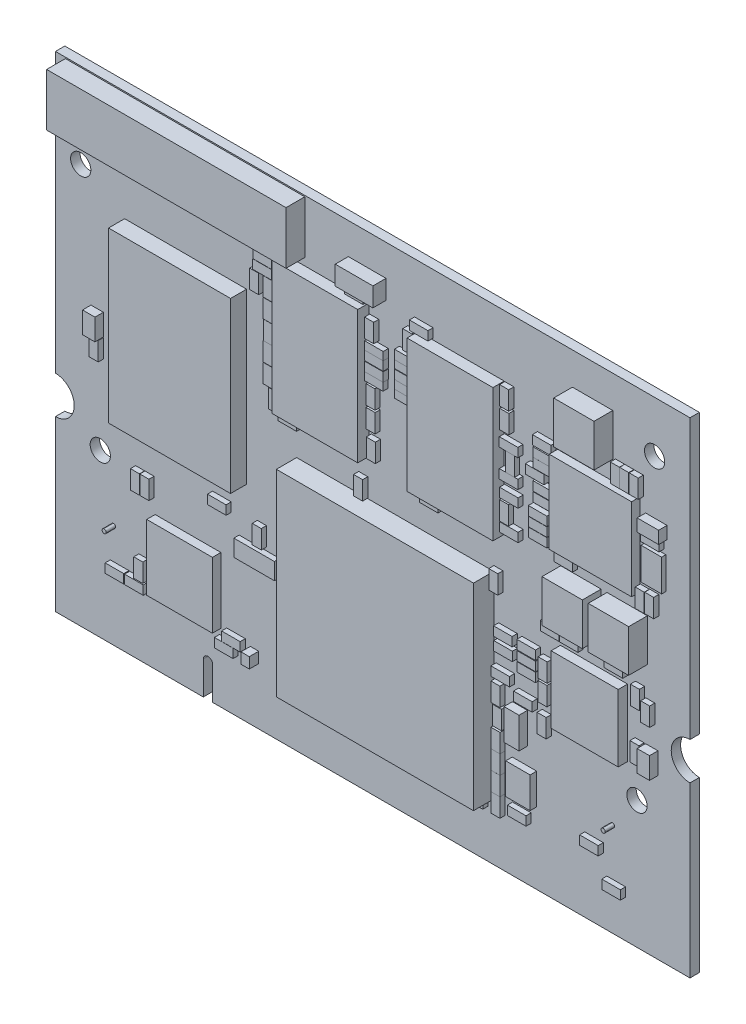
SolidWorks part; units mm, degrees
ref_plane "Front Plane" through (0, 0, 0) normal (0, 0, 1) x (1, 0, 0)
ref_plane "Top Plane" through (0, 0, 0) normal (0, 1, 0) x (1, 0, 0)
ref_plane "Right Plane" through (0, 0, 0) normal (1, 0, 0) x (0, 0, -1)
sketch "Sketch1" plane through (0, 0, 0) normal (0, 0, 1) x (1, 0, 0)
  line L0 (75.2145, 18.001) -> (75.2145, 0)
  line L1 (75.2145, 0) -> (24.3637, 0)
  line L2 (24.3637, 0) -> (24.3637, 3.5001)
  line L3 (23.3655, 3.5001) -> (23.3655, 0)
  line L4 (23.3655, 0) -> (7.6149, 0)
  line L5 (7.6149, 0) -> (7.6149, 18.001)
  line L6 (7.6149, 21.9989) -> (7.6149, 51.689)
  line L7 (7.6149, 51.689) -> (75.2145, 51.689)
  line L8 (75.2145, 51.689) -> (75.2145, 21.9989)
  arc A0 (75.2145, 21.9989) -> (73.2155, 20) centre (75.2145, 20) ccw
  arc A1 (73.2155, 20) -> (75.2145, 18.001) centre (75.2145, 20) ccw
  arc A2 (24.3637, 3.5001) -> (23.8658, 4.0005) centre (23.8646, 3.5014) ccw
  arc A3 (23.8658, 4.0005) -> (23.3655, 3.5001) centre (23.8658, 3.5001) ccw
  arc A4 (7.6149, 18.001) -> (9.6139, 20) centre (7.6149, 20) ccw
  arc A5 (9.6139, 20) -> (7.6149, 21.9989) centre (7.6149, 20) ccw
extrude "BOARD" add sketch "Sketch1" along normal blind 1 separate body
ref_plane "Plane1" through (0, 0, 1.0008) normal (0, 0, 1) x (1, 0, 0)
sketch "Sketch2" plane through (0, 0, 1.0008) normal (0, 0, 1) x (1, 0, 0)
  line L0 (56.2818, 10.921) -> (58.8818, 10.921)
  line L1 (58.8818, 10.921) -> (58.8818, 7.621)
  line L2 (58.8818, 7.621) -> (56.2818, 7.621)
  line L3 (56.2818, 7.621) -> (56.2818, 10.921)
extrude "NX3225SA-1" add sketch "Sketch2" along normal blind 0.7 separate body
sketch "Sketch3" plane through (0, 0, 1.0008) normal (0, 0, 1) x (1, 0, 0)
  line L0 (28.3794, 7.1755) -> (28.3794, 6.0325)
  line L1 (28.3794, 6.0325) -> (29.2684, 6.0325)
  line L2 (29.2684, 6.0325) -> (29.2684, 7.1755)
  line L3 (29.2684, 7.1755) -> (28.3794, 7.1755)
extrude "PVQFN_16N-1" add sketch "Sketch3" along normal blind 1 separate body
sketch "Sketch4" plane through (0, 0, 0) normal (0, 0, 1) x (1, 0, 0)
  line L0 (8.3744, 39.6824) -> (8.3744, 36.3804)
  line L1 (8.3744, 36.3804) -> (10.6604, 36.3804)
  line L2 (10.6604, 36.3804) -> (10.6604, 39.6824)
  line L3 (10.6604, 39.6824) -> (8.3744, 39.6824)
extrude "SC-70-6-1" add sketch "Sketch4" against normal blind 1.0998 separate body
sketch "Sketch10" plane through (0, 0, 0) normal (0, 0, 1) x (1, 0, 0)
  line L0 (70.4466, 37.7706) -> (72.6468, 37.7706)
  line L1 (72.6468, 37.7706) -> (72.6468, 34.3705)
  line L2 (72.6468, 34.3705) -> (70.4466, 34.3705)
  line L3 (70.4466, 34.3705) -> (70.4466, 37.7706)
extrude "MLP2012S1R0T-1" add sketch "Sketch10" along normal blind 1.4501 separate body
sketch "Sketch11" plane through (0, 0, 0) normal (0, 0, 1) x (1, 0, 0)
  line L0 (42.7759, 11.1399) -> (42.7759, 11.242)
  line L1 (42.7759, 11.242) -> (42.7609, 11.242)
  line L2 (42.7609, 11.242) -> (42.7609, 11.872)
  line L3 (42.7609, 11.872) -> (42.7759, 11.872)
  line L4 (42.7759, 11.872) -> (42.7759, 11.9741)
  line L5 (42.7759, 11.9741) -> (43.0761, 11.9741)
  line L6 (43.0761, 11.9741) -> (43.0761, 11.872)
  line L7 (43.0761, 11.872) -> (43.0911, 11.872)
  line L8 (43.0911, 11.872) -> (43.0911, 11.242)
  line L9 (43.0911, 11.242) -> (43.0761, 11.242)
  line L10 (43.0761, 11.242) -> (43.0761, 11.1399)
  line L11 (43.0761, 11.1399) -> (42.7759, 11.1399)
extrude "0201_CC-1" add sketch "Sketch11" against normal blind 0.3299 separate body
sketch "Sketch12" plane through (0, 0, 0) normal (0, 0, 1) x (1, 0, 0)
  line L0 (42.5811, 18.1125) -> (42.479, 18.1125)
  line L1 (42.479, 18.1125) -> (42.479, 18.0975)
  line L2 (42.479, 18.0975) -> (41.849, 18.0975)
  line L3 (41.849, 18.0975) -> (41.849, 18.1125)
  line L4 (41.849, 18.1125) -> (41.7469, 18.1125)
  line L5 (41.7469, 18.1125) -> (41.7469, 18.4127)
  line L6 (41.7469, 18.4127) -> (41.849, 18.4127)
  line L7 (41.849, 18.4127) -> (41.849, 18.4277)
  line L8 (41.849, 18.4277) -> (42.479, 18.4277)
  line L9 (42.479, 18.4277) -> (42.479, 18.4127)
  line L10 (42.479, 18.4127) -> (42.5811, 18.4127)
  line L11 (42.5811, 18.4127) -> (42.5811, 18.1125)
extrude "0201_CC-2" add sketch "Sketch12" against normal blind 0.3299 separate body
sketch "Sketch13" plane through (0, 0, 0) normal (0, 0, 1) x (1, 0, 0)
  line L0 (42.5473, 14.9499) -> (42.5473, 15.052)
  line L1 (42.5473, 15.052) -> (42.5323, 15.052)
  line L2 (42.5323, 15.052) -> (42.5323, 15.682)
  line L3 (42.5323, 15.682) -> (42.5473, 15.682)
  line L4 (42.5473, 15.682) -> (42.5473, 15.7841)
  line L5 (42.5473, 15.7841) -> (42.8475, 15.7841)
  line L6 (42.8475, 15.7841) -> (42.8475, 15.682)
  line L7 (42.8475, 15.682) -> (42.8625, 15.682)
  line L8 (42.8625, 15.682) -> (42.8625, 15.052)
  line L9 (42.8625, 15.052) -> (42.8475, 15.052)
  line L10 (42.8475, 15.052) -> (42.8475, 14.9499)
  line L11 (42.8475, 14.9499) -> (42.5473, 14.9499)
extrude "0201_CC-3" add sketch "Sketch13" against normal blind 0.3299 separate body
sketch "Sketch14" plane through (0, 0, 0) normal (0, 0, 1) x (1, 0, 0)
  line L0 (40.6761, 17.2489) -> (40.574, 17.2489)
  line L1 (40.574, 17.2489) -> (40.574, 17.2339)
  line L2 (40.574, 17.2339) -> (39.944, 17.2339)
  line L3 (39.944, 17.2339) -> (39.944, 17.2489)
  line L4 (39.944, 17.2489) -> (39.8419, 17.2489)
  line L5 (39.8419, 17.2489) -> (39.8419, 17.5491)
  line L6 (39.8419, 17.5491) -> (39.944, 17.5491)
  line L7 (39.944, 17.5491) -> (39.944, 17.5641)
  line L8 (39.944, 17.5641) -> (40.574, 17.5641)
  line L9 (40.574, 17.5641) -> (40.574, 17.5491)
  line L10 (40.574, 17.5491) -> (40.6761, 17.5491)
  line L11 (40.6761, 17.5491) -> (40.6761, 17.2489)
extrude "0201_CC-4" add sketch "Sketch14" against normal blind 0.3299 separate body
sketch "Sketch15" plane through (0, 0, 0) normal (0, 0, 1) x (1, 0, 0)
  line L0 (41.9331, 15.7841) -> (41.9331, 15.682)
  line L1 (41.9331, 15.682) -> (41.9481, 15.682)
  line L2 (41.9481, 15.682) -> (41.9481, 15.052)
  line L3 (41.9481, 15.052) -> (41.9331, 15.052)
  line L4 (41.9331, 15.052) -> (41.9331, 14.9499)
  line L5 (41.9331, 14.9499) -> (41.6329, 14.9499)
  line L6 (41.6329, 14.9499) -> (41.6329, 15.052)
  line L7 (41.6329, 15.052) -> (41.6179, 15.052)
  line L8 (41.6179, 15.052) -> (41.6179, 15.682)
  line L9 (41.6179, 15.682) -> (41.6329, 15.682)
  line L10 (41.6329, 15.682) -> (41.6329, 15.7841)
  line L11 (41.6329, 15.7841) -> (41.9331, 15.7841)
extrude "0201_CC-5" add sketch "Sketch15" against normal blind 0.3299 separate body
sketch "Sketch16" plane through (0, 0, 0) normal (0, 0, 1) x (1, 0, 0)
  line L0 (41.7469, 14.2217) -> (41.849, 14.2217)
  line L1 (41.849, 14.2217) -> (41.849, 14.2367)
  line L2 (41.849, 14.2367) -> (42.479, 14.2367)
  line L3 (42.479, 14.2367) -> (42.479, 14.2217)
  line L4 (42.479, 14.2217) -> (42.5811, 14.2217)
  line L5 (42.5811, 14.2217) -> (42.5811, 13.9215)
  line L6 (42.5811, 13.9215) -> (42.479, 13.9215)
  line L7 (42.479, 13.9215) -> (42.479, 13.9065)
  line L8 (42.479, 13.9065) -> (41.849, 13.9065)
  line L9 (41.849, 13.9065) -> (41.849, 13.9215)
  line L10 (41.849, 13.9215) -> (41.7469, 13.9215)
  line L11 (41.7469, 13.9215) -> (41.7469, 14.2217)
extrude "0201_CC-6" add sketch "Sketch16" against normal blind 0.3299 separate body
sketch "Sketch17" plane through (0, 0, 0) normal (0, 0, 1) x (1, 0, 0)
  line L0 (46.7383, 11.7495) -> (46.7383, 11.8516)
  line L1 (46.7383, 11.8516) -> (46.7233, 11.8516)
  line L2 (46.7233, 11.8516) -> (46.7233, 12.4816)
  line L3 (46.7233, 12.4816) -> (46.7383, 12.4816)
  line L4 (46.7383, 12.4816) -> (46.7383, 12.5837)
  line L5 (46.7383, 12.5837) -> (47.0385, 12.5837)
  line L6 (47.0385, 12.5837) -> (47.0385, 12.4816)
  line L7 (47.0385, 12.4816) -> (47.0535, 12.4816)
  line L8 (47.0535, 12.4816) -> (47.0535, 11.8516)
  line L9 (47.0535, 11.8516) -> (47.0385, 11.8516)
  line L10 (47.0385, 11.8516) -> (47.0385, 11.7495)
  line L11 (47.0385, 11.7495) -> (46.7383, 11.7495)
extrude "0201_CC-7" add sketch "Sketch17" against normal blind 0.3299 separate body
sketch "Sketch18" plane through (0, 0, 0) normal (0, 0, 1) x (1, 0, 0)
  line L0 (49.0581, 16.5123) -> (48.956, 16.5123)
  line L1 (48.956, 16.5123) -> (48.956, 16.4973)
  line L2 (48.956, 16.4973) -> (48.326, 16.4973)
  line L3 (48.326, 16.4973) -> (48.326, 16.5123)
  line L4 (48.326, 16.5123) -> (48.2239, 16.5123)
  line L5 (48.2239, 16.5123) -> (48.2239, 16.8125)
  line L6 (48.2239, 16.8125) -> (48.326, 16.8125)
  line L7 (48.326, 16.8125) -> (48.326, 16.8275)
  line L8 (48.326, 16.8275) -> (48.956, 16.8275)
  line L9 (48.956, 16.8275) -> (48.956, 16.8125)
  line L10 (48.956, 16.8125) -> (49.0581, 16.8125)
  line L11 (49.0581, 16.8125) -> (49.0581, 16.5123)
extrude "0201_CC-8" add sketch "Sketch18" against normal blind 0.3299 separate body
sketch "Sketch19" plane through (0, 0, 0) normal (0, 0, 1) x (1, 0, 0)
  line L0 (49.3121, 17.1219) -> (49.21, 17.1219)
  line L1 (49.21, 17.1219) -> (49.21, 17.1069)
  line L2 (49.21, 17.1069) -> (48.58, 17.1069)
  line L3 (48.58, 17.1069) -> (48.58, 17.1219)
  line L4 (48.58, 17.1219) -> (48.4779, 17.1219)
  line L5 (48.4779, 17.1219) -> (48.4779, 17.4221)
  line L6 (48.4779, 17.4221) -> (48.58, 17.4221)
  line L7 (48.58, 17.4221) -> (48.58, 17.4371)
  line L8 (48.58, 17.4371) -> (49.21, 17.4371)
  line L9 (49.21, 17.4371) -> (49.21, 17.4221)
  line L10 (49.21, 17.4221) -> (49.3121, 17.4221)
  line L11 (49.3121, 17.4221) -> (49.3121, 17.1219)
extrude "0201_CC-9" add sketch "Sketch19" against normal blind 0.3299 separate body
sketch "Sketch20" plane through (0, 0, 0) normal (0, 0, 1) x (1, 0, 0)
  line L0 (42.1409, 20.5379) -> (42.1409, 20.64)
  line L1 (42.1409, 20.64) -> (42.1259, 20.64)
  line L2 (42.1259, 20.64) -> (42.1259, 21.27)
  line L3 (42.1259, 21.27) -> (42.1409, 21.27)
  line L4 (42.1409, 21.27) -> (42.1409, 21.3721)
  line L5 (42.1409, 21.3721) -> (42.4411, 21.3721)
  line L6 (42.4411, 21.3721) -> (42.4411, 21.27)
  line L7 (42.4411, 21.27) -> (42.4561, 21.27)
  line L8 (42.4561, 21.27) -> (42.4561, 20.64)
  line L9 (42.4561, 20.64) -> (42.4411, 20.64)
  line L10 (42.4411, 20.64) -> (42.4411, 20.5379)
  line L11 (42.4411, 20.5379) -> (42.1409, 20.5379)
extrude "0201_CC-10" add sketch "Sketch20" against normal blind 0.3299 separate body
sketch "Sketch21" plane through (0, 0, 0) normal (0, 0, 1) x (1, 0, 0)
  line L0 (40.4899, 20.5379) -> (40.4899, 20.64)
  line L1 (40.4899, 20.64) -> (40.4749, 20.64)
  line L2 (40.4749, 20.64) -> (40.4749, 21.27)
  line L3 (40.4749, 21.27) -> (40.4899, 21.27)
  line L4 (40.4899, 21.27) -> (40.4899, 21.3721)
  line L5 (40.4899, 21.3721) -> (40.7901, 21.3721)
  line L6 (40.7901, 21.3721) -> (40.7901, 21.27)
  line L7 (40.7901, 21.27) -> (40.8051, 21.27)
  line L8 (40.8051, 21.27) -> (40.8051, 20.64)
  line L9 (40.8051, 20.64) -> (40.7901, 20.64)
  line L10 (40.7901, 20.64) -> (40.7901, 20.5379)
  line L11 (40.7901, 20.5379) -> (40.4899, 20.5379)
extrude "0201_CC-11" add sketch "Sketch21" against normal blind 0.3299 separate body
sketch "Sketch22" plane through (0, 0, 0) normal (0, 0, 1) x (1, 0, 0)
  line L0 (46.9539, 21.1051) -> (47.056, 21.1051)
  line L1 (47.056, 21.1051) -> (47.056, 21.1201)
  line L2 (47.056, 21.1201) -> (47.686, 21.1201)
  line L3 (47.686, 21.1201) -> (47.686, 21.1051)
  line L4 (47.686, 21.1051) -> (47.7881, 21.1051)
  line L5 (47.7881, 21.1051) -> (47.7881, 20.8049)
  line L6 (47.7881, 20.8049) -> (47.686, 20.8049)
  line L7 (47.686, 20.8049) -> (47.686, 20.7899)
  line L8 (47.686, 20.7899) -> (47.056, 20.7899)
  line L9 (47.056, 20.7899) -> (47.056, 20.8049)
  line L10 (47.056, 20.8049) -> (46.9539, 20.8049)
  line L11 (46.9539, 20.8049) -> (46.9539, 21.1051)
extrude "0201_CC-12" add sketch "Sketch22" against normal blind 0.3299 separate body
sketch "Sketch23" plane through (0, 0, 0) normal (0, 0, 1) x (1, 0, 0)
  line L0 (41.1249, 20.5379) -> (41.1249, 20.64)
  line L1 (41.1249, 20.64) -> (41.1099, 20.64)
  line L2 (41.1099, 20.64) -> (41.1099, 21.27)
  line L3 (41.1099, 21.27) -> (41.1249, 21.27)
  line L4 (41.1249, 21.27) -> (41.1249, 21.3721)
  line L5 (41.1249, 21.3721) -> (41.4251, 21.3721)
  line L6 (41.4251, 21.3721) -> (41.4251, 21.27)
  line L7 (41.4251, 21.27) -> (41.4401, 21.27)
  line L8 (41.4401, 21.27) -> (41.4401, 20.64)
  line L9 (41.4401, 20.64) -> (41.4251, 20.64)
  line L10 (41.4251, 20.64) -> (41.4251, 20.5379)
  line L11 (41.4251, 20.5379) -> (41.1249, 20.5379)
extrude "0201_CC-13" add sketch "Sketch23" against normal blind 0.3299 separate body
sketch "Sketch24" plane through (0, 0, 0) normal (0, 0, 1) x (1, 0, 0)
  line L0 (43.7789, 21.3591) -> (43.881, 21.3591)
  line L1 (43.881, 21.3591) -> (43.881, 21.3741)
  line L2 (43.881, 21.3741) -> (44.511, 21.3741)
  line L3 (44.511, 21.3741) -> (44.511, 21.3591)
  line L4 (44.511, 21.3591) -> (44.6131, 21.3591)
  line L5 (44.6131, 21.3591) -> (44.6131, 21.0589)
  line L6 (44.6131, 21.0589) -> (44.511, 21.0589)
  line L7 (44.511, 21.0589) -> (44.511, 21.0439)
  line L8 (44.511, 21.0439) -> (43.881, 21.0439)
  line L9 (43.881, 21.0439) -> (43.881, 21.0589)
  line L10 (43.881, 21.0589) -> (43.7789, 21.0589)
  line L11 (43.7789, 21.0589) -> (43.7789, 21.3591)
extrude "0201_CC-14" add sketch "Sketch24" against normal blind 0.3299 separate body
sketch "Sketch25" plane through (0, 0, 0) normal (0, 0, 1) x (1, 0, 0)
  line L0 (45.4299, 21.3591) -> (45.532, 21.3591)
  line L1 (45.532, 21.3591) -> (45.532, 21.3741)
  line L2 (45.532, 21.3741) -> (46.162, 21.3741)
  line L3 (46.162, 21.3741) -> (46.162, 21.3591)
  line L4 (46.162, 21.3591) -> (46.2641, 21.3591)
  line L5 (46.2641, 21.3591) -> (46.2641, 21.0589)
  line L6 (46.2641, 21.0589) -> (46.162, 21.0589)
  line L7 (46.162, 21.0589) -> (46.162, 21.0439)
  line L8 (46.162, 21.0439) -> (45.532, 21.0439)
  line L9 (45.532, 21.0439) -> (45.532, 21.0589)
  line L10 (45.532, 21.0589) -> (45.4299, 21.0589)
  line L11 (45.4299, 21.0589) -> (45.4299, 21.3591)
extrude "0201_CC-15" add sketch "Sketch25" against normal blind 0.3299 separate body
sketch "Sketch26" plane through (0, 0, 0) normal (0, 0, 1) x (1, 0, 0)
  line L0 (40.6631, 19.7211) -> (40.6631, 19.619)
  line L1 (40.6631, 19.619) -> (40.6781, 19.619)
  line L2 (40.6781, 19.619) -> (40.6781, 18.989)
  line L3 (40.6781, 18.989) -> (40.6631, 18.989)
  line L4 (40.6631, 18.989) -> (40.6631, 18.8869)
  line L5 (40.6631, 18.8869) -> (40.3629, 18.8869)
  line L6 (40.3629, 18.8869) -> (40.3629, 18.989)
  line L7 (40.3629, 18.989) -> (40.3479, 18.989)
  line L8 (40.3479, 18.989) -> (40.3479, 19.619)
  line L9 (40.3479, 19.619) -> (40.3629, 19.619)
  line L10 (40.3629, 19.619) -> (40.3629, 19.7211)
  line L11 (40.3629, 19.7211) -> (40.6631, 19.7211)
extrude "0201_CC-16" add sketch "Sketch26" against normal blind 0.3299 separate body
sketch "Sketch27" plane through (0, 0, 0) normal (0, 0, 1) x (1, 0, 0)
  line L0 (39.8419, 18.2349) -> (39.944, 18.2349)
  line L1 (39.944, 18.2349) -> (39.944, 18.2499)
  line L2 (39.944, 18.2499) -> (40.574, 18.2499)
  line L3 (40.574, 18.2499) -> (40.574, 18.2349)
  line L4 (40.574, 18.2349) -> (40.6761, 18.2349)
  line L5 (40.6761, 18.2349) -> (40.6761, 17.9347)
  line L6 (40.6761, 17.9347) -> (40.574, 17.9347)
  line L7 (40.574, 17.9347) -> (40.574, 17.9197)
  line L8 (40.574, 17.9197) -> (39.944, 17.9197)
  line L9 (39.944, 17.9197) -> (39.944, 17.9347)
  line L10 (39.944, 17.9347) -> (39.8419, 17.9347)
  line L11 (39.8419, 17.9347) -> (39.8419, 18.2349)
extrude "0201_CC-17" add sketch "Sketch27" against normal blind 0.3299 separate body
sketch "Sketch28" plane through (0, 0, 0) normal (0, 0, 1) x (1, 0, 0)
  line L0 (41.4381, 13.9469) -> (41.336, 13.9469)
  line L1 (41.336, 13.9469) -> (41.336, 13.9319)
  line L2 (41.336, 13.9319) -> (40.706, 13.9319)
  line L3 (40.706, 13.9319) -> (40.706, 13.9469)
  line L4 (40.706, 13.9469) -> (40.6039, 13.9469)
  line L5 (40.6039, 13.9469) -> (40.6039, 14.2471)
  line L6 (40.6039, 14.2471) -> (40.706, 14.2471)
  line L7 (40.706, 14.2471) -> (40.706, 14.2621)
  line L8 (40.706, 14.2621) -> (41.336, 14.2621)
  line L9 (41.336, 14.2621) -> (41.336, 14.2471)
  line L10 (41.336, 14.2471) -> (41.4381, 14.2471)
  line L11 (41.4381, 14.2471) -> (41.4381, 13.9469)
extrude "0201_CC-18" add sketch "Sketch28" against normal blind 0.3299 separate body
sketch "Sketch29" plane through (0, 0, 0) normal (0, 0, 1) x (1, 0, 0)
  line L0 (40.9047, 12.2959) -> (40.8026, 12.2959)
  line L1 (40.8026, 12.2959) -> (40.8026, 12.2809)
  line L2 (40.8026, 12.2809) -> (40.1726, 12.2809)
  line L3 (40.1726, 12.2809) -> (40.1726, 12.2959)
  line L4 (40.1726, 12.2959) -> (40.0705, 12.2959)
  line L5 (40.0705, 12.2959) -> (40.0705, 12.5961)
  line L6 (40.0705, 12.5961) -> (40.1726, 12.5961)
  line L7 (40.1726, 12.5961) -> (40.1726, 12.6111)
  line L8 (40.1726, 12.6111) -> (40.8026, 12.6111)
  line L9 (40.8026, 12.6111) -> (40.8026, 12.5961)
  line L10 (40.8026, 12.5961) -> (40.9047, 12.5961)
  line L11 (40.9047, 12.5961) -> (40.9047, 12.2959)
extrude "0201_CC-19" add sketch "Sketch29" against normal blind 0.3299 separate body
sketch "Sketch30" plane through (0, 0, 0) normal (0, 0, 1) x (1, 0, 0)
  line L0 (46.9669, 13.4259) -> (46.9669, 13.528)
  line L1 (46.9669, 13.528) -> (46.9519, 13.528)
  line L2 (46.9519, 13.528) -> (46.9519, 14.158)
  line L3 (46.9519, 14.158) -> (46.9669, 14.158)
  line L4 (46.9669, 14.158) -> (46.9669, 14.2601)
  line L5 (46.9669, 14.2601) -> (47.2671, 14.2601)
  line L6 (47.2671, 14.2601) -> (47.2671, 14.158)
  line L7 (47.2671, 14.158) -> (47.2821, 14.158)
  line L8 (47.2821, 14.158) -> (47.2821, 13.528)
  line L9 (47.2821, 13.528) -> (47.2671, 13.528)
  line L10 (47.2671, 13.528) -> (47.2671, 13.4259)
  line L11 (47.2671, 13.4259) -> (46.9669, 13.4259)
extrude "0201_CC-20" add sketch "Sketch30" against normal blind 0.3299 separate body
sketch "Sketch31" plane through (0, 0, 0) normal (0, 0, 1) x (1, 0, 0)
  line L0 (40.6761, 16.2329) -> (40.574, 16.2329)
  line L1 (40.574, 16.2329) -> (40.574, 16.2179)
  line L2 (40.574, 16.2179) -> (39.944, 16.2179)
  line L3 (39.944, 16.2179) -> (39.944, 16.2329)
  line L4 (39.944, 16.2329) -> (39.8419, 16.2329)
  line L5 (39.8419, 16.2329) -> (39.8419, 16.5331)
  line L6 (39.8419, 16.5331) -> (39.944, 16.5331)
  line L7 (39.944, 16.5331) -> (39.944, 16.5481)
  line L8 (39.944, 16.5481) -> (40.574, 16.5481)
  line L9 (40.574, 16.5481) -> (40.574, 16.5331)
  line L10 (40.574, 16.5331) -> (40.6761, 16.5331)
  line L11 (40.6761, 16.5331) -> (40.6761, 16.2329)
extrude "0201_CC-21" add sketch "Sketch31" against normal blind 0.3299 separate body
sketch "Sketch32" plane through (0, 0, 0) normal (0, 0, 1) x (1, 0, 0)
  line L0 (38.4579, 15.7119) -> (38.4579, 15.814)
  line L1 (38.4579, 15.814) -> (38.4429, 15.814)
  line L2 (38.4429, 15.814) -> (38.4429, 16.444)
  line L3 (38.4429, 16.444) -> (38.4579, 16.444)
  line L4 (38.4579, 16.444) -> (38.4579, 16.5461)
  line L5 (38.4579, 16.5461) -> (38.7581, 16.5461)
  line L6 (38.7581, 16.5461) -> (38.7581, 16.444)
  line L7 (38.7581, 16.444) -> (38.7731, 16.444)
  line L8 (38.7731, 16.444) -> (38.7731, 15.814)
  line L9 (38.7731, 15.814) -> (38.7581, 15.814)
  line L10 (38.7581, 15.814) -> (38.7581, 15.7119)
  line L11 (38.7581, 15.7119) -> (38.4579, 15.7119)
extrude "0201_CC-22" add sketch "Sketch32" against normal blind 0.3299 separate body
sketch "Sketch33" plane through (0, 0, 0) normal (0, 0, 1) x (1, 0, 0)
  line L0 (47.7667, 12.2913) -> (47.8688, 12.2913)
  line L1 (47.8688, 12.2913) -> (47.8688, 12.3063)
  line L2 (47.8688, 12.3063) -> (48.4988, 12.3063)
  line L3 (48.4988, 12.3063) -> (48.4988, 12.2913)
  line L4 (48.4988, 12.2913) -> (48.6009, 12.2913)
  line L5 (48.6009, 12.2913) -> (48.6009, 11.9911)
  line L6 (48.6009, 11.9911) -> (48.4988, 11.9911)
  line L7 (48.4988, 11.9911) -> (48.4988, 11.9761)
  line L8 (48.4988, 11.9761) -> (47.8688, 11.9761)
  line L9 (47.8688, 11.9761) -> (47.8688, 11.9911)
  line L10 (47.8688, 11.9911) -> (47.7667, 11.9911)
  line L11 (47.7667, 11.9911) -> (47.7667, 12.2913)
extrude "0201_CC-23" add sketch "Sketch33" against normal blind 0.3299 separate body
sketch "Sketch34" plane through (0, 0, 0) normal (0, 0, 1) x (1, 0, 0)
  line L0 (47.0301, 13.0787) -> (47.1322, 13.0787)
  line L1 (47.1322, 13.0787) -> (47.1322, 13.0937)
  line L2 (47.1322, 13.0937) -> (47.7622, 13.0937)
  line L3 (47.7622, 13.0937) -> (47.7622, 13.0787)
  line L4 (47.7622, 13.0787) -> (47.8643, 13.0787)
  line L5 (47.8643, 13.0787) -> (47.8643, 12.7785)
  line L6 (47.8643, 12.7785) -> (47.7622, 12.7785)
  line L7 (47.7622, 12.7785) -> (47.7622, 12.7635)
  line L8 (47.7622, 12.7635) -> (47.1322, 12.7635)
  line L9 (47.1322, 12.7635) -> (47.1322, 12.7785)
  line L10 (47.1322, 12.7785) -> (47.0301, 12.7785)
  line L11 (47.0301, 12.7785) -> (47.0301, 13.0787)
extrude "0201_CC-24" add sketch "Sketch34" against normal blind 0.3299 separate body
sketch "Sketch35" plane through (0, 0, 0) normal (0, 0, 1) x (1, 0, 0)
  line L0 (41.3789, 11.7749) -> (41.3789, 11.877)
  line L1 (41.3789, 11.877) -> (41.3639, 11.877)
  line L2 (41.3639, 11.877) -> (41.3639, 12.507)
  line L3 (41.3639, 12.507) -> (41.3789, 12.507)
  line L4 (41.3789, 12.507) -> (41.3789, 12.6091)
  line L5 (41.3789, 12.6091) -> (41.6791, 12.6091)
  line L6 (41.6791, 12.6091) -> (41.6791, 12.507)
  line L7 (41.6791, 12.507) -> (41.6941, 12.507)
  line L8 (41.6941, 12.507) -> (41.6941, 11.877)
  line L9 (41.6941, 11.877) -> (41.6791, 11.877)
  line L10 (41.6791, 11.877) -> (41.6791, 11.7749)
  line L11 (41.6791, 11.7749) -> (41.3789, 11.7749)
extrude "0201_CC-25" add sketch "Sketch35" against normal blind 0.3299 separate body
sketch "Sketch36" plane through (0, 0, 0) normal (0, 0, 1) x (1, 0, 0)
  line L0 (39.4609, 14.2217) -> (39.563, 14.2217)
  line L1 (39.563, 14.2217) -> (39.563, 14.2367)
  line L2 (39.563, 14.2367) -> (40.193, 14.2367)
  line L3 (40.193, 14.2367) -> (40.193, 14.2217)
  line L4 (40.193, 14.2217) -> (40.2951, 14.2217)
  line L5 (40.2951, 14.2217) -> (40.2951, 13.9215)
  line L6 (40.2951, 13.9215) -> (40.193, 13.9215)
  line L7 (40.193, 13.9215) -> (40.193, 13.9065)
  line L8 (40.193, 13.9065) -> (39.563, 13.9065)
  line L9 (39.563, 13.9065) -> (39.563, 13.9215)
  line L10 (39.563, 13.9215) -> (39.4609, 13.9215)
  line L11 (39.4609, 13.9215) -> (39.4609, 14.2217)
extrude "0201_CC-26" add sketch "Sketch36" against normal blind 0.3299 separate body
sketch "Sketch37" plane through (0, 0, 0) normal (0, 0, 1) x (1, 0, 0)
  line L0 (48.6049, 9.6751) -> (48.707, 9.6751)
  line L1 (48.707, 9.6751) -> (48.707, 9.6901)
  line L2 (48.707, 9.6901) -> (49.337, 9.6901)
  line L3 (49.337, 9.6901) -> (49.337, 9.6751)
  line L4 (49.337, 9.6751) -> (49.4391, 9.6751)
  line L5 (49.4391, 9.6751) -> (49.4391, 9.3749)
  line L6 (49.4391, 9.3749) -> (49.337, 9.3749)
  line L7 (49.337, 9.3749) -> (49.337, 9.3599)
  line L8 (49.337, 9.3599) -> (48.707, 9.3599)
  line L9 (48.707, 9.3599) -> (48.707, 9.3749)
  line L10 (48.707, 9.3749) -> (48.6049, 9.3749)
  line L11 (48.6049, 9.3749) -> (48.6049, 9.6751)
extrude "0201_CC-27" add sketch "Sketch37" against normal blind 0.3299 separate body
sketch "Sketch38" plane through (0, 0, 0) normal (0, 0, 1) x (1, 0, 0)
  line L0 (45.8239, 11.7495) -> (45.8239, 11.8516)
  line L1 (45.8239, 11.8516) -> (45.8089, 11.8516)
  line L2 (45.8089, 11.8516) -> (45.8089, 12.4816)
  line L3 (45.8089, 12.4816) -> (45.8239, 12.4816)
  line L4 (45.8239, 12.4816) -> (45.8239, 12.5837)
  line L5 (45.8239, 12.5837) -> (46.1241, 12.5837)
  line L6 (46.1241, 12.5837) -> (46.1241, 12.4816)
  line L7 (46.1241, 12.4816) -> (46.1391, 12.4816)
  line L8 (46.1391, 12.4816) -> (46.1391, 11.8516)
  line L9 (46.1391, 11.8516) -> (46.1241, 11.8516)
  line L10 (46.1241, 11.8516) -> (46.1241, 11.7495)
  line L11 (46.1241, 11.7495) -> (45.8239, 11.7495)
extrude "0201_CC-28" add sketch "Sketch38" against normal blind 0.3299 separate body
sketch "Sketch39" plane through (0, 0, 0) normal (0, 0, 1) x (1, 0, 0)
  line L0 (38.2501, 18.1209) -> (38.2501, 18.0188)
  line L1 (38.2501, 18.0188) -> (38.2651, 18.0188)
  line L2 (38.2651, 18.0188) -> (38.2651, 17.3888)
  line L3 (38.2651, 17.3888) -> (38.2501, 17.3888)
  line L4 (38.2501, 17.3888) -> (38.2501, 17.2867)
  line L5 (38.2501, 17.2867) -> (37.9499, 17.2867)
  line L6 (37.9499, 17.2867) -> (37.9499, 17.3888)
  line L7 (37.9499, 17.3888) -> (37.9349, 17.3888)
  line L8 (37.9349, 17.3888) -> (37.9349, 18.0188)
  line L9 (37.9349, 18.0188) -> (37.9499, 18.0188)
  line L10 (37.9499, 18.0188) -> (37.9499, 18.1209)
  line L11 (37.9499, 18.1209) -> (38.2501, 18.1209)
extrude "0201_CC-29" add sketch "Sketch39" against normal blind 0.3299 separate body
sketch "Sketch40" plane through (0, 0, 0) normal (0, 0, 1) x (1, 0, 0)
  line L0 (45.8109, 17.6761) -> (45.913, 17.6761)
  line L1 (45.913, 17.6761) -> (45.913, 17.6911)
  line L2 (45.913, 17.6911) -> (46.543, 17.6911)
  line L3 (46.543, 17.6911) -> (46.543, 17.6761)
  line L4 (46.543, 17.6761) -> (46.6451, 17.6761)
  line L5 (46.6451, 17.6761) -> (46.6451, 17.3759)
  line L6 (46.6451, 17.3759) -> (46.543, 17.3759)
  line L7 (46.543, 17.3759) -> (46.543, 17.3609)
  line L8 (46.543, 17.3609) -> (45.913, 17.3609)
  line L9 (45.913, 17.3609) -> (45.913, 17.3759)
  line L10 (45.913, 17.3759) -> (45.8109, 17.3759)
  line L11 (45.8109, 17.3759) -> (45.8109, 17.6761)
extrude "0201_CC-30" add sketch "Sketch40" against normal blind 0.3299 separate body
sketch "Sketch41" plane through (0, 0, 0) normal (0, 0, 1) x (1, 0, 0)
  line L0 (46.7591, 15.7841) -> (46.7591, 15.682)
  line L1 (46.7591, 15.682) -> (46.7741, 15.682)
  line L2 (46.7741, 15.682) -> (46.7741, 15.052)
  line L3 (46.7741, 15.052) -> (46.7591, 15.052)
  line L4 (46.7591, 15.052) -> (46.7591, 14.9499)
  line L5 (46.7591, 14.9499) -> (46.4589, 14.9499)
  line L6 (46.4589, 14.9499) -> (46.4589, 15.052)
  line L7 (46.4589, 15.052) -> (46.4439, 15.052)
  line L8 (46.4439, 15.052) -> (46.4439, 15.682)
  line L9 (46.4439, 15.682) -> (46.4589, 15.682)
  line L10 (46.4589, 15.682) -> (46.4589, 15.7841)
  line L11 (46.4589, 15.7841) -> (46.7591, 15.7841)
extrude "0201_CC-31" add sketch "Sketch41" against normal blind 0.3299 separate body
sketch "Sketch42" plane through (0, 0, 0) normal (0, 0, 1) x (1, 0, 0)
  line L0 (47.5973, 15.7841) -> (47.5973, 15.682)
  line L1 (47.5973, 15.682) -> (47.6123, 15.682)
  line L2 (47.6123, 15.682) -> (47.6123, 15.052)
  line L3 (47.6123, 15.052) -> (47.5973, 15.052)
  line L4 (47.5973, 15.052) -> (47.5973, 14.9499)
  line L5 (47.5973, 14.9499) -> (47.2971, 14.9499)
  line L6 (47.2971, 14.9499) -> (47.2971, 15.052)
  line L7 (47.2971, 15.052) -> (47.2821, 15.052)
  line L8 (47.2821, 15.052) -> (47.2821, 15.682)
  line L9 (47.2821, 15.682) -> (47.2971, 15.682)
  line L10 (47.2971, 15.682) -> (47.2971, 15.7841)
  line L11 (47.2971, 15.7841) -> (47.5973, 15.7841)
extrude "0201_CC-32" add sketch "Sketch42" against normal blind 0.3299 separate body
sketch "Sketch43" plane through (0, 0, 0) normal (0, 0, 1) x (1, 0, 0)
  line L0 (46.3149, 13.2865) -> (46.2128, 13.2865)
  line L1 (46.2128, 13.2865) -> (46.2128, 13.2715)
  line L2 (46.2128, 13.2715) -> (45.5828, 13.2715)
  line L3 (45.5828, 13.2715) -> (45.5828, 13.2865)
  line L4 (45.5828, 13.2865) -> (45.4807, 13.2865)
  line L5 (45.4807, 13.2865) -> (45.4807, 13.5867)
  line L6 (45.4807, 13.5867) -> (45.5828, 13.5867)
  line L7 (45.5828, 13.5867) -> (45.5828, 13.6017)
  line L8 (45.5828, 13.6017) -> (46.2128, 13.6017)
  line L9 (46.2128, 13.6017) -> (46.2128, 13.5867)
  line L10 (46.2128, 13.5867) -> (46.3149, 13.5867)
  line L11 (46.3149, 13.5867) -> (46.3149, 13.2865)
extrude "0201_CC-33" add sketch "Sketch43" against normal blind 0.3299 separate body
sketch "Sketch44" plane through (0, 0, 0) normal (0, 0, 1) x (1, 0, 0)
  line L0 (45.4807, 14.2217) -> (45.5828, 14.2217)
  line L1 (45.5828, 14.2217) -> (45.5828, 14.2367)
  line L2 (45.5828, 14.2367) -> (46.2128, 14.2367)
  line L3 (46.2128, 14.2367) -> (46.2128, 14.2217)
  line L4 (46.2128, 14.2217) -> (46.3149, 14.2217)
  line L5 (46.3149, 14.2217) -> (46.3149, 13.9215)
  line L6 (46.3149, 13.9215) -> (46.2128, 13.9215)
  line L7 (46.2128, 13.9215) -> (46.2128, 13.9065)
  line L8 (46.2128, 13.9065) -> (45.5828, 13.9065)
  line L9 (45.5828, 13.9065) -> (45.5828, 13.9215)
  line L10 (45.5828, 13.9215) -> (45.4807, 13.9215)
  line L11 (45.4807, 13.9215) -> (45.4807, 14.2217)
extrude "0201_CC-34" add sketch "Sketch44" against normal blind 0.3299 separate body
sketch "Sketch45" plane through (0, 0, 0) normal (0, 0, 1) x (1, 0, 0)
  line L0 (41.7469, 19.0223) -> (41.849, 19.0223)
  line L1 (41.849, 19.0223) -> (41.849, 19.0373)
  line L2 (41.849, 19.0373) -> (42.479, 19.0373)
  line L3 (42.479, 19.0373) -> (42.479, 19.0223)
  line L4 (42.479, 19.0223) -> (42.5811, 19.0223)
  line L5 (42.5811, 19.0223) -> (42.5811, 18.7221)
  line L6 (42.5811, 18.7221) -> (42.479, 18.7221)
  line L7 (42.479, 18.7221) -> (42.479, 18.7071)
  line L8 (42.479, 18.7071) -> (41.849, 18.7071)
  line L9 (41.849, 18.7071) -> (41.849, 18.7221)
  line L10 (41.849, 18.7221) -> (41.7469, 18.7221)
  line L11 (41.7469, 18.7221) -> (41.7469, 19.0223)
extrude "0201_CC-35" add sketch "Sketch45" against normal blind 0.3299 separate body
sketch "Sketch46" plane through (0, 0, 0) normal (0, 0, 1) x (1, 0, 0)
  line L0 (47.6905, 14.1709) -> (47.7926, 14.1709)
  line L1 (47.7926, 14.1709) -> (47.7926, 14.1859)
  line L2 (47.7926, 14.1859) -> (48.4226, 14.1859)
  line L3 (48.4226, 14.1859) -> (48.4226, 14.1709)
  line L4 (48.4226, 14.1709) -> (48.5247, 14.1709)
  line L5 (48.5247, 14.1709) -> (48.5247, 13.8707)
  line L6 (48.5247, 13.8707) -> (48.4226, 13.8707)
  line L7 (48.4226, 13.8707) -> (48.4226, 13.8557)
  line L8 (48.4226, 13.8557) -> (47.7926, 13.8557)
  line L9 (47.7926, 13.8557) -> (47.7926, 13.8707)
  line L10 (47.7926, 13.8707) -> (47.6905, 13.8707)
  line L11 (47.6905, 13.8707) -> (47.6905, 14.1709)
extrude "0201_CC-36" add sketch "Sketch46" against normal blind 0.3299 separate body
sketch "Sketch47" plane through (0, 0, 0) normal (0, 0, 1) x (1, 0, 0)
  line L0 (47.3349, 17.4221) -> (47.437, 17.4221)
  line L1 (47.437, 17.4221) -> (47.437, 17.4371)
  line L2 (47.437, 17.4371) -> (48.067, 17.4371)
  line L3 (48.067, 17.4371) -> (48.067, 17.4221)
  line L4 (48.067, 17.4221) -> (48.1691, 17.4221)
  line L5 (48.1691, 17.4221) -> (48.1691, 17.1219)
  line L6 (48.1691, 17.1219) -> (48.067, 17.1219)
  line L7 (48.067, 17.1219) -> (48.067, 17.1069)
  line L8 (48.067, 17.1069) -> (47.437, 17.1069)
  line L9 (47.437, 17.1069) -> (47.437, 17.1219)
  line L10 (47.437, 17.1219) -> (47.3349, 17.1219)
  line L11 (47.3349, 17.1219) -> (47.3349, 17.4221)
extrude "0201_CC-37" add sketch "Sketch47" against normal blind 0.3299 separate body
sketch "Sketch48" plane through (0, 0, 0) normal (0, 0, 1) x (1, 0, 0)
  line L0 (43.7789, 13.4089) -> (43.881, 13.4089)
  line L1 (43.881, 13.4089) -> (43.881, 13.4239)
  line L2 (43.881, 13.4239) -> (44.511, 13.4239)
  line L3 (44.511, 13.4239) -> (44.511, 13.4089)
  line L4 (44.511, 13.4089) -> (44.6131, 13.4089)
  line L5 (44.6131, 13.4089) -> (44.6131, 13.1087)
  line L6 (44.6131, 13.1087) -> (44.511, 13.1087)
  line L7 (44.511, 13.1087) -> (44.511, 13.0937)
  line L8 (44.511, 13.0937) -> (43.881, 13.0937)
  line L9 (43.881, 13.0937) -> (43.881, 13.1087)
  line L10 (43.881, 13.1087) -> (43.7789, 13.1087)
  line L11 (43.7789, 13.1087) -> (43.7789, 13.4089)
extrude "0201_CC-38" add sketch "Sketch48" against normal blind 0.3299 separate body
sketch "Sketch49" plane through (0, 0, 0) normal (0, 0, 1) x (1, 0, 0)
  line L0 (43.7789, 12.7231) -> (43.881, 12.7231)
  line L1 (43.881, 12.7231) -> (43.881, 12.7381)
  line L2 (43.881, 12.7381) -> (44.511, 12.7381)
  line L3 (44.511, 12.7381) -> (44.511, 12.7231)
  line L4 (44.511, 12.7231) -> (44.6131, 12.7231)
  line L5 (44.6131, 12.7231) -> (44.6131, 12.4229)
  line L6 (44.6131, 12.4229) -> (44.511, 12.4229)
  line L7 (44.511, 12.4229) -> (44.511, 12.4079)
  line L8 (44.511, 12.4079) -> (43.881, 12.4079)
  line L9 (43.881, 12.4079) -> (43.881, 12.4229)
  line L10 (43.881, 12.4229) -> (43.7789, 12.4229)
  line L11 (43.7789, 12.4229) -> (43.7789, 12.7231)
extrude "0201_CC-39" add sketch "Sketch49" against normal blind 0.3299 separate body
sketch "Sketch50" plane through (0, 0, 0) normal (0, 0, 1) x (1, 0, 0)
  line L0 (42.1787, 17.1427) -> (42.2808, 17.1427)
  line L1 (42.2808, 17.1427) -> (42.2808, 17.1577)
  line L2 (42.2808, 17.1577) -> (42.9108, 17.1577)
  line L3 (42.9108, 17.1577) -> (42.9108, 17.1427)
  line L4 (42.9108, 17.1427) -> (43.0129, 17.1427)
  line L5 (43.0129, 17.1427) -> (43.0129, 16.8425)
  line L6 (43.0129, 16.8425) -> (42.9108, 16.8425)
  line L7 (42.9108, 16.8425) -> (42.9108, 16.8275)
  line L8 (42.9108, 16.8275) -> (42.2808, 16.8275)
  line L9 (42.2808, 16.8275) -> (42.2808, 16.8425)
  line L10 (42.2808, 16.8425) -> (42.1787, 16.8425)
  line L11 (42.1787, 16.8425) -> (42.1787, 17.1427)
extrude "0201_CC-40" add sketch "Sketch50" against normal blind 0.3299 separate body
sketch "Sketch51" plane through (0, 0, 0) normal (0, 0, 1) x (1, 0, 0)
  line L0 (43.8511, 14.1755) -> (43.749, 14.1755)
  line L1 (43.749, 14.1755) -> (43.749, 14.1605)
  line L2 (43.749, 14.1605) -> (43.119, 14.1605)
  line L3 (43.119, 14.1605) -> (43.119, 14.1755)
  line L4 (43.119, 14.1755) -> (43.0169, 14.1755)
  line L5 (43.0169, 14.1755) -> (43.0169, 14.4757)
  line L6 (43.0169, 14.4757) -> (43.119, 14.4757)
  line L7 (43.119, 14.4757) -> (43.119, 14.4907)
  line L8 (43.119, 14.4907) -> (43.749, 14.4907)
  line L9 (43.749, 14.4907) -> (43.749, 14.4757)
  line L10 (43.749, 14.4757) -> (43.8511, 14.4757)
  line L11 (43.8511, 14.4757) -> (43.8511, 14.1755)
extrude "0201_CC-41" add sketch "Sketch51" against normal blind 0.3299 separate body
sketch "Sketch52" plane through (0, 0, 0) normal (0, 0, 1) x (1, 0, 0)
  line L0 (47.4619, 19.0223) -> (47.564, 19.0223)
  line L1 (47.564, 19.0223) -> (47.564, 19.0373)
  line L2 (47.564, 19.0373) -> (48.194, 19.0373)
  line L3 (48.194, 19.0373) -> (48.194, 19.0223)
  line L4 (48.194, 19.0223) -> (48.2961, 19.0223)
  line L5 (48.2961, 19.0223) -> (48.2961, 18.7221)
  line L6 (48.2961, 18.7221) -> (48.194, 18.7221)
  line L7 (48.194, 18.7221) -> (48.194, 18.7071)
  line L8 (48.194, 18.7071) -> (47.564, 18.7071)
  line L9 (47.564, 18.7071) -> (47.564, 18.7221)
  line L10 (47.564, 18.7221) -> (47.4619, 18.7221)
  line L11 (47.4619, 18.7221) -> (47.4619, 19.0223)
extrude "0201_CC-42" add sketch "Sketch52" against normal blind 0.3299 separate body
sketch "Sketch53" plane through (0, 0, 0) normal (0, 0, 1) x (1, 0, 0)
  line L0 (39.3931, 18.0701) -> (39.3931, 17.968)
  line L1 (39.3931, 17.968) -> (39.4081, 17.968)
  line L2 (39.4081, 17.968) -> (39.4081, 17.338)
  line L3 (39.4081, 17.338) -> (39.3931, 17.338)
  line L4 (39.3931, 17.338) -> (39.3931, 17.2359)
  line L5 (39.3931, 17.2359) -> (39.0929, 17.2359)
  line L6 (39.0929, 17.2359) -> (39.0929, 17.338)
  line L7 (39.0929, 17.338) -> (39.0779, 17.338)
  line L8 (39.0779, 17.338) -> (39.0779, 17.968)
  line L9 (39.0779, 17.968) -> (39.0929, 17.968)
  line L10 (39.0929, 17.968) -> (39.0929, 18.0701)
  line L11 (39.0929, 18.0701) -> (39.3931, 18.0701)
extrude "0201_CC-43" add sketch "Sketch53" against normal blind 0.3299 separate body
sketch "Sketch54" plane through (0, 0, 0) normal (0, 0, 1) x (1, 0, 0)
  line L0 (43.0761, 20.6101) -> (43.0761, 20.508)
  line L1 (43.0761, 20.508) -> (43.0911, 20.508)
  line L2 (43.0911, 20.508) -> (43.0911, 19.878)
  line L3 (43.0911, 19.878) -> (43.0761, 19.878)
  line L4 (43.0761, 19.878) -> (43.0761, 19.7759)
  line L5 (43.0761, 19.7759) -> (42.7759, 19.7759)
  line L6 (42.7759, 19.7759) -> (42.7759, 19.878)
  line L7 (42.7759, 19.878) -> (42.7609, 19.878)
  line L8 (42.7609, 19.878) -> (42.7609, 20.508)
  line L9 (42.7609, 20.508) -> (42.7759, 20.508)
  line L10 (42.7759, 20.508) -> (42.7759, 20.6101)
  line L11 (42.7759, 20.6101) -> (43.0761, 20.6101)
extrude "0201_CC-44" add sketch "Sketch54" against normal blind 0.3299 separate body
sketch "Sketch55" plane through (0, 0, 0) normal (0, 0, 1) x (1, 0, 0)
  line L0 (42.1409, 11.7749) -> (42.1409, 11.877)
  line L1 (42.1409, 11.877) -> (42.1259, 11.877)
  line L2 (42.1259, 11.877) -> (42.1259, 12.507)
  line L3 (42.1259, 12.507) -> (42.1409, 12.507)
  line L4 (42.1409, 12.507) -> (42.1409, 12.6091)
  line L5 (42.1409, 12.6091) -> (42.4411, 12.6091)
  line L6 (42.4411, 12.6091) -> (42.4411, 12.507)
  line L7 (42.4411, 12.507) -> (42.4561, 12.507)
  line L8 (42.4561, 12.507) -> (42.4561, 11.877)
  line L9 (42.4561, 11.877) -> (42.4411, 11.877)
  line L10 (42.4411, 11.877) -> (42.4411, 11.7749)
  line L11 (42.4411, 11.7749) -> (42.1409, 11.7749)
extrude "0201_CC-45" add sketch "Sketch55" against normal blind 0.3299 separate body
sketch "Sketch56" plane through (0, 0, 0) normal (0, 0, 1) x (1, 0, 0)
  line L0 (43.0891, 13.3119) -> (42.987, 13.3119)
  line L1 (42.987, 13.3119) -> (42.987, 13.2969)
  line L2 (42.987, 13.2969) -> (42.357, 13.2969)
  line L3 (42.357, 13.2969) -> (42.357, 13.3119)
  line L4 (42.357, 13.3119) -> (42.2549, 13.3119)
  line L5 (42.2549, 13.3119) -> (42.2549, 13.6121)
  line L6 (42.2549, 13.6121) -> (42.357, 13.6121)
  line L7 (42.357, 13.6121) -> (42.357, 13.6271)
  line L8 (42.357, 13.6271) -> (42.987, 13.6271)
  line L9 (42.987, 13.6271) -> (42.987, 13.6121)
  line L10 (42.987, 13.6121) -> (43.0891, 13.6121)
  line L11 (43.0891, 13.6121) -> (43.0891, 13.3119)
extrude "0201_CC-46" add sketch "Sketch56" against normal blind 0.3299 separate body
sketch "Sketch57" plane through (0, 0, 0) normal (0, 0, 1) x (1, 0, 0)
  line L0 (49.3873, 10.9985) -> (49.4894, 10.9985)
  line L1 (49.4894, 10.9985) -> (49.4894, 11.0134)
  line L2 (49.4894, 11.0134) -> (50.1193, 11.0134)
  line L3 (50.1193, 11.0134) -> (50.1193, 10.9985)
  line L4 (50.1193, 10.9985) -> (50.2214, 10.9985)
  line L5 (50.2214, 10.9985) -> (50.2214, 10.6982)
  line L6 (50.2214, 10.6982) -> (50.1193, 10.6982)
  line L7 (50.1193, 10.6982) -> (50.1193, 10.6832)
  line L8 (50.1193, 10.6832) -> (49.4894, 10.6832)
  line L9 (49.4894, 10.6832) -> (49.4894, 10.6982)
  line L10 (49.4894, 10.6982) -> (49.3873, 10.6982)
  line L11 (49.3873, 10.6982) -> (49.3873, 10.9985)
extrude "0201_CC-47" add sketch "Sketch57" against normal blind 0.3299 separate body
sketch "Sketch58" plane through (0, 0, 0) normal (0, 0, 1) x (1, 0, 0)
  line L0 (46.9539, 20.3431) -> (47.056, 20.3431)
  line L1 (47.056, 20.3431) -> (47.056, 20.3581)
  line L2 (47.056, 20.3581) -> (47.686, 20.3581)
  line L3 (47.686, 20.3581) -> (47.686, 20.3431)
  line L4 (47.686, 20.3431) -> (47.7881, 20.3431)
  line L5 (47.7881, 20.3431) -> (47.7881, 20.0429)
  line L6 (47.7881, 20.0429) -> (47.686, 20.0429)
  line L7 (47.686, 20.0429) -> (47.686, 20.0279)
  line L8 (47.686, 20.0279) -> (47.056, 20.0279)
  line L9 (47.056, 20.0279) -> (47.056, 20.0429)
  line L10 (47.056, 20.0429) -> (46.9539, 20.0429)
  line L11 (46.9539, 20.0429) -> (46.9539, 20.3431)
extrude "0201_CC-48" add sketch "Sketch58" against normal blind 0.3299 separate body
sketch "Sketch59" plane through (0, 0, 0) normal (0, 0, 1) x (1, 0, 0)
  line L0 (48.5821, 21.1346) -> (48.6842, 21.1346)
  line L1 (48.6842, 21.1346) -> (48.6842, 21.1496)
  line L2 (48.6842, 21.1496) -> (49.3141, 21.1496)
  line L3 (49.3141, 21.1496) -> (49.3141, 21.1346)
  line L4 (49.3141, 21.1346) -> (49.4162, 21.1346)
  line L5 (49.4162, 21.1346) -> (49.4162, 20.8344)
  line L6 (49.4162, 20.8344) -> (49.3141, 20.8344)
  line L7 (49.3141, 20.8344) -> (49.3141, 20.8194)
  line L8 (49.3141, 20.8194) -> (48.6842, 20.8194)
  line L9 (48.6842, 20.8194) -> (48.6842, 20.8344)
  line L10 (48.6842, 20.8344) -> (48.5821, 20.8344)
  line L11 (48.5821, 20.8344) -> (48.5821, 21.1346)
extrude "0201_CC-49" add sketch "Sketch59" against normal blind 0.3299 separate body
sketch "Sketch60" plane through (0, 0, 0) normal (0, 0, 1) x (1, 0, 0)
  line L0 (43.7241, 18.7221) -> (43.622, 18.7221)
  line L1 (43.622, 18.7221) -> (43.622, 18.7071)
  line L2 (43.622, 18.7071) -> (42.992, 18.7071)
  line L3 (42.992, 18.7071) -> (42.992, 18.7221)
  line L4 (42.992, 18.7221) -> (42.8899, 18.7221)
  line L5 (42.8899, 18.7221) -> (42.8899, 19.0223)
  line L6 (42.8899, 19.0223) -> (42.992, 19.0223)
  line L7 (42.992, 19.0223) -> (42.992, 19.0373)
  line L8 (42.992, 19.0373) -> (43.622, 19.0373)
  line L9 (43.622, 19.0373) -> (43.622, 19.0223)
  line L10 (43.622, 19.0223) -> (43.7241, 19.0223)
  line L11 (43.7241, 19.0223) -> (43.7241, 18.7221)
extrude "0201_CC-50" add sketch "Sketch60" against normal blind 0.3299 separate body
sketch "Sketch61" plane through (0, 0, 0) normal (0, 0, 1) x (1, 0, 0)
  line L0 (45.0619, 11.7495) -> (45.0619, 11.8516)
  line L1 (45.0619, 11.8516) -> (45.0469, 11.8516)
  line L2 (45.0469, 11.8516) -> (45.0469, 12.4816)
  line L3 (45.0469, 12.4816) -> (45.0619, 12.4816)
  line L4 (45.0619, 12.4816) -> (45.0619, 12.5837)
  line L5 (45.0619, 12.5837) -> (45.3621, 12.5837)
  line L6 (45.3621, 12.5837) -> (45.3621, 12.4816)
  line L7 (45.3621, 12.4816) -> (45.3771, 12.4816)
  line L8 (45.3771, 12.4816) -> (45.3771, 11.8516)
  line L9 (45.3771, 11.8516) -> (45.3621, 11.8516)
  line L10 (45.3621, 11.8516) -> (45.3621, 11.7495)
  line L11 (45.3621, 11.7495) -> (45.0619, 11.7495)
extrude "0201_CC-51" add sketch "Sketch61" against normal blind 0.3299 separate body
sketch "Sketch62" plane through (0, 0, 0) normal (0, 0, 1) x (1, 0, 0)
  line L0 (44.6639, 16.3091) -> (44.5618, 16.3091)
  line L1 (44.5618, 16.3091) -> (44.5618, 16.2941)
  line L2 (44.5618, 16.2941) -> (43.9318, 16.2941)
  line L3 (43.9318, 16.2941) -> (43.9318, 16.3091)
  line L4 (43.9318, 16.3091) -> (43.8297, 16.3091)
  line L5 (43.8297, 16.3091) -> (43.8297, 16.6093)
  line L6 (43.8297, 16.6093) -> (43.9318, 16.6093)
  line L7 (43.9318, 16.6093) -> (43.9318, 16.6243)
  line L8 (43.9318, 16.6243) -> (44.5618, 16.6243)
  line L9 (44.5618, 16.6243) -> (44.5618, 16.6093)
  line L10 (44.5618, 16.6093) -> (44.6639, 16.6093)
  line L11 (44.6639, 16.6093) -> (44.6639, 16.3091)
extrude "0201_CC-52" add sketch "Sketch62" against normal blind 0.3299 separate body
sketch "Sketch63" plane through (0, 0, 0) normal (0, 0, 1) x (1, 0, 0)
  line L0 (47.8125, 10.9985) -> (47.9146, 10.9985)
  line L1 (47.9146, 10.9985) -> (47.9146, 11.0134)
  line L2 (47.9146, 11.0134) -> (48.5445, 11.0134)
  line L3 (48.5445, 11.0134) -> (48.5445, 10.9985)
  line L4 (48.5445, 10.9985) -> (48.6466, 10.9985)
  line L5 (48.6466, 10.9985) -> (48.6466, 10.6982)
  line L6 (48.6466, 10.6982) -> (48.5445, 10.6982)
  line L7 (48.5445, 10.6982) -> (48.5445, 10.6832)
  line L8 (48.5445, 10.6832) -> (47.9146, 10.6832)
  line L9 (47.9146, 10.6832) -> (47.9146, 10.6982)
  line L10 (47.9146, 10.6982) -> (47.8125, 10.6982)
  line L11 (47.8125, 10.6982) -> (47.8125, 10.9985)
extrude "0201_CC-53" add sketch "Sketch63" against normal blind 0.3299 separate body
sketch "Sketch64" plane through (0, 0, 0) normal (0, 0, 1) x (1, 0, 0)
  line L0 (39.7871, 11.4069) -> (39.685, 11.4069)
  line L1 (39.685, 11.4069) -> (39.685, 11.3919)
  line L2 (39.685, 11.3919) -> (39.055, 11.3919)
  line L3 (39.055, 11.3919) -> (39.055, 11.4069)
  line L4 (39.055, 11.4069) -> (38.9529, 11.4069)
  line L5 (38.9529, 11.4069) -> (38.9529, 11.7071)
  line L6 (38.9529, 11.7071) -> (39.055, 11.7071)
  line L7 (39.055, 11.7071) -> (39.055, 11.7221)
  line L8 (39.055, 11.7221) -> (39.685, 11.7221)
  line L9 (39.685, 11.7221) -> (39.685, 11.7071)
  line L10 (39.685, 11.7071) -> (39.7871, 11.7071)
  line L11 (39.7871, 11.7071) -> (39.7871, 11.4069)
extrude "0201_CC-54" add sketch "Sketch64" against normal blind 0.3299 separate body
sketch "Sketch65" plane through (0, 0, 0) normal (0, 0, 1) x (1, 0, 0)
  line L0 (49.8625, 9.4889) -> (49.8625, 9.591)
  line L1 (49.8625, 9.591) -> (49.8475, 9.591)
  line L2 (49.8475, 9.591) -> (49.8475, 10.221)
  line L3 (49.8475, 10.221) -> (49.8625, 10.221)
  line L4 (49.8625, 10.221) -> (49.8625, 10.3231)
  line L5 (49.8625, 10.3231) -> (50.1627, 10.3231)
  line L6 (50.1627, 10.3231) -> (50.1627, 10.221)
  line L7 (50.1627, 10.221) -> (50.1777, 10.221)
  line L8 (50.1777, 10.221) -> (50.1777, 9.591)
  line L9 (50.1777, 9.591) -> (50.1627, 9.591)
  line L10 (50.1627, 9.591) -> (50.1627, 9.4889)
  line L11 (50.1627, 9.4889) -> (49.8625, 9.4889)
extrude "0201_CC-55" add sketch "Sketch65" against normal blind 0.3299 separate body
sketch "Sketch66" plane through (0, 0, 0) normal (0, 0, 1) x (1, 0, 0)
  line L0 (46.1386, 8.5971) -> (46.1386, 8.495)
  line L1 (46.1386, 8.495) -> (46.1536, 8.495)
  line L2 (46.1536, 8.495) -> (46.1536, 7.8651)
  line L3 (46.1536, 7.8651) -> (46.1386, 7.8651)
  line L4 (46.1386, 7.8651) -> (46.1386, 7.763)
  line L5 (46.1386, 7.763) -> (45.8384, 7.763)
  line L6 (45.8384, 7.763) -> (45.8384, 7.8651)
  line L7 (45.8384, 7.8651) -> (45.8234, 7.8651)
  line L8 (45.8234, 7.8651) -> (45.8234, 8.495)
  line L9 (45.8234, 8.495) -> (45.8384, 8.495)
  line L10 (45.8384, 8.495) -> (45.8384, 8.5971)
  line L11 (45.8384, 8.5971) -> (46.1386, 8.5971)
extrude "0201_CC-56" add sketch "Sketch66" against normal blind 0.3299 separate body
sketch "Sketch67" plane through (0, 0, 0) normal (0, 0, 1) x (1, 0, 0)
  line L0 (47.752, 8.5387) -> (47.8541, 8.5387)
  line L1 (47.8541, 8.5387) -> (47.8541, 8.5537)
  line L2 (47.8541, 8.5537) -> (48.484, 8.5537)
  line L3 (48.484, 8.5537) -> (48.484, 8.5387)
  line L4 (48.484, 8.5387) -> (48.5861, 8.5387)
  line L5 (48.5861, 8.5387) -> (48.5861, 8.2385)
  line L6 (48.5861, 8.2385) -> (48.484, 8.2385)
  line L7 (48.484, 8.2385) -> (48.484, 8.2235)
  line L8 (48.484, 8.2235) -> (47.8541, 8.2235)
  line L9 (47.8541, 8.2235) -> (47.8541, 8.2385)
  line L10 (47.8541, 8.2385) -> (47.752, 8.2385)
  line L11 (47.752, 8.2385) -> (47.752, 8.5387)
extrude "0201_CC-57" add sketch "Sketch67" against normal blind 0.3299 separate body
sketch "Sketch68" plane through (0, 0, 0) normal (0, 0, 1) x (1, 0, 0)
  line L0 (43.7789, 12.0119) -> (43.881, 12.0119)
  line L1 (43.881, 12.0119) -> (43.881, 12.0269)
  line L2 (43.881, 12.0269) -> (44.511, 12.0269)
  line L3 (44.511, 12.0269) -> (44.511, 12.0119)
  line L4 (44.511, 12.0119) -> (44.6131, 12.0119)
  line L5 (44.6131, 12.0119) -> (44.6131, 11.7117)
  line L6 (44.6131, 11.7117) -> (44.511, 11.7117)
  line L7 (44.511, 11.7117) -> (44.511, 11.6967)
  line L8 (44.511, 11.6967) -> (43.881, 11.6967)
  line L9 (43.881, 11.6967) -> (43.881, 11.7117)
  line L10 (43.881, 11.7117) -> (43.7789, 11.7117)
  line L11 (43.7789, 11.7117) -> (43.7789, 12.0119)
extrude "0201_CC-58" add sketch "Sketch68" against normal blind 0.3299 separate body
sketch "Sketch69" plane through (0, 0, 0) normal (0, 0, 1) x (1, 0, 0)
  line L0 (49.3873, 14.9609) -> (49.4894, 14.9609)
  line L1 (49.4894, 14.9609) -> (49.4894, 14.9758)
  line L2 (49.4894, 14.9758) -> (50.1193, 14.9758)
  line L3 (50.1193, 14.9758) -> (50.1193, 14.9609)
  line L4 (50.1193, 14.9609) -> (50.2214, 14.9609)
  line L5 (50.2214, 14.9609) -> (50.2214, 14.6606)
  line L6 (50.2214, 14.6606) -> (50.1193, 14.6606)
  line L7 (50.1193, 14.6606) -> (50.1193, 14.6456)
  line L8 (50.1193, 14.6456) -> (49.4894, 14.6456)
  line L9 (49.4894, 14.6456) -> (49.4894, 14.6606)
  line L10 (49.4894, 14.6606) -> (49.3873, 14.6606)
  line L11 (49.3873, 14.6606) -> (49.3873, 14.9609)
extrude "0201_CC-59" add sketch "Sketch69" against normal blind 0.3299 separate body
sketch "Sketch70" plane through (0, 0, 0) normal (0, 0, 1) x (1, 0, 0)
  line L0 (48.8719, 12.5369) -> (48.8719, 12.639)
  line L1 (48.8719, 12.639) -> (48.8569, 12.639)
  line L2 (48.8569, 12.639) -> (48.8569, 13.269)
  line L3 (48.8569, 13.269) -> (48.8719, 13.269)
  line L4 (48.8719, 13.269) -> (48.8719, 13.3711)
  line L5 (48.8719, 13.3711) -> (49.1721, 13.3711)
  line L6 (49.1721, 13.3711) -> (49.1721, 13.269)
  line L7 (49.1721, 13.269) -> (49.1871, 13.269)
  line L8 (49.1871, 13.269) -> (49.1871, 12.639)
  line L9 (49.1871, 12.639) -> (49.1721, 12.639)
  line L10 (49.1721, 12.639) -> (49.1721, 12.5369)
  line L11 (49.1721, 12.5369) -> (48.8719, 12.5369)
extrude "0201_CC-60" add sketch "Sketch70" against normal blind 0.3299 separate body
sketch "Sketch71" plane through (0, 0, 0) normal (0, 0, 1) x (1, 0, 0)
  line L0 (43.7789, 17.6761) -> (43.881, 17.6761)
  line L1 (43.881, 17.6761) -> (43.881, 17.6911)
  line L2 (43.881, 17.6911) -> (44.511, 17.6911)
  line L3 (44.511, 17.6911) -> (44.511, 17.6761)
  line L4 (44.511, 17.6761) -> (44.6131, 17.6761)
  line L5 (44.6131, 17.6761) -> (44.6131, 17.3759)
  line L6 (44.6131, 17.3759) -> (44.511, 17.3759)
  line L7 (44.511, 17.3759) -> (44.511, 17.3609)
  line L8 (44.511, 17.3609) -> (43.881, 17.3609)
  line L9 (43.881, 17.3609) -> (43.881, 17.3759)
  line L10 (43.881, 17.3759) -> (43.7789, 17.3759)
  line L11 (43.7789, 17.3759) -> (43.7789, 17.6761)
extrude "0201_CC-61" add sketch "Sketch71" against normal blind 0.3299 separate body
sketch "Sketch72" plane through (0, 0, 0) normal (0, 0, 1) x (1, 0, 0)
  line L0 (47.4619, 18.4127) -> (47.564, 18.4127)
  line L1 (47.564, 18.4127) -> (47.564, 18.4277)
  line L2 (47.564, 18.4277) -> (48.194, 18.4277)
  line L3 (48.194, 18.4277) -> (48.194, 18.4127)
  line L4 (48.194, 18.4127) -> (48.2961, 18.4127)
  line L5 (48.2961, 18.4127) -> (48.2961, 18.1125)
  line L6 (48.2961, 18.1125) -> (48.194, 18.1125)
  line L7 (48.194, 18.1125) -> (48.194, 18.0975)
  line L8 (48.194, 18.0975) -> (47.564, 18.0975)
  line L9 (47.564, 18.0975) -> (47.564, 18.1125)
  line L10 (47.564, 18.1125) -> (47.4619, 18.1125)
  line L11 (47.4619, 18.1125) -> (47.4619, 18.4127)
extrude "0201_CC-62" add sketch "Sketch72" against normal blind 0.3299 separate body
sketch "Sketch73" plane through (0, 0, 0) normal (0, 0, 1) x (1, 0, 0)
  line L0 (48.4101, 15.7841) -> (48.4101, 15.682)
  line L1 (48.4101, 15.682) -> (48.4251, 15.682)
  line L2 (48.4251, 15.682) -> (48.4251, 15.052)
  line L3 (48.4251, 15.052) -> (48.4101, 15.052)
  line L4 (48.4101, 15.052) -> (48.4101, 14.9499)
  line L5 (48.4101, 14.9499) -> (48.1099, 14.9499)
  line L6 (48.1099, 14.9499) -> (48.1099, 15.052)
  line L7 (48.1099, 15.052) -> (48.0949, 15.052)
  line L8 (48.0949, 15.052) -> (48.0949, 15.682)
  line L9 (48.0949, 15.682) -> (48.1099, 15.682)
  line L10 (48.1099, 15.682) -> (48.1099, 15.7841)
  line L11 (48.1099, 15.7841) -> (48.4101, 15.7841)
extrude "0201_CC-63" add sketch "Sketch73" against normal blind 0.3299 separate body
sketch "Sketch74" plane through (0, 0, 0) normal (0, 0, 1) x (1, 0, 0)
  line L0 (49.4386, 14.4206) -> (49.5407, 14.4206)
  line L1 (49.5407, 14.4206) -> (49.5407, 14.4356)
  line L2 (49.5407, 14.4356) -> (50.1706, 14.4356)
  line L3 (50.1706, 14.4356) -> (50.1706, 14.4206)
  line L4 (50.1706, 14.4206) -> (50.2727, 14.4206)
  line L5 (50.2727, 14.4206) -> (50.2727, 14.1204)
  line L6 (50.2727, 14.1204) -> (50.1706, 14.1204)
  line L7 (50.1706, 14.1204) -> (50.1706, 14.1054)
  line L8 (50.1706, 14.1054) -> (49.5407, 14.1054)
  line L9 (49.5407, 14.1054) -> (49.5407, 14.1204)
  line L10 (49.5407, 14.1204) -> (49.4386, 14.1204)
  line L11 (49.4386, 14.1204) -> (49.4386, 14.4206)
extrude "0201_CC-64" add sketch "Sketch74" against normal blind 0.3299 separate body
sketch "Sketch75" plane through (0, 0, 0) normal (0, 0, 1) x (1, 0, 0)
  line L0 (43.4571, 16.6223) -> (43.4571, 16.5202)
  line L1 (43.4571, 16.5202) -> (43.4721, 16.5202)
  line L2 (43.4721, 16.5202) -> (43.4721, 15.8902)
  line L3 (43.4721, 15.8902) -> (43.4571, 15.8902)
  line L4 (43.4571, 15.8902) -> (43.4571, 15.7881)
  line L5 (43.4571, 15.7881) -> (43.1569, 15.7881)
  line L6 (43.1569, 15.7881) -> (43.1569, 15.8902)
  line L7 (43.1569, 15.8902) -> (43.1419, 15.8902)
  line L8 (43.1419, 15.8902) -> (43.1419, 16.5202)
  line L9 (43.1419, 16.5202) -> (43.1569, 16.5202)
  line L10 (43.1569, 16.5202) -> (43.1569, 16.6223)
  line L11 (43.1569, 16.6223) -> (43.4571, 16.6223)
extrude "0201_CC-65" add sketch "Sketch75" against normal blind 0.3299 separate body
sketch "Sketch76" plane through (0, 0, 0) normal (0, 0, 1) x (1, 0, 0)
  line L0 (41.4381, 13.3119) -> (41.336, 13.3119)
  line L1 (41.336, 13.3119) -> (41.336, 13.2969)
  line L2 (41.336, 13.2969) -> (40.706, 13.2969)
  line L3 (40.706, 13.2969) -> (40.706, 13.3119)
  line L4 (40.706, 13.3119) -> (40.6039, 13.3119)
  line L5 (40.6039, 13.3119) -> (40.6039, 13.6121)
  line L6 (40.6039, 13.6121) -> (40.706, 13.6121)
  line L7 (40.706, 13.6121) -> (40.706, 13.6271)
  line L8 (40.706, 13.6271) -> (41.336, 13.6271)
  line L9 (41.336, 13.6271) -> (41.336, 13.6121)
  line L10 (41.336, 13.6121) -> (41.4381, 13.6121)
  line L11 (41.4381, 13.6121) -> (41.4381, 13.3119)
extrude "0201_CC-66" add sketch "Sketch76" against normal blind 0.3299 separate body
sketch "Sketch78" plane through (0, 0, 1.0008) normal (0, 0, 1) x (1, 0, 0)
  circle A0 centre (71.4451, 46.2559) radius 1.0795
sketch "Sketch79" plane through (0, 0, 1.0008) normal (0, 0, 1) x (1, 0, 0)
  circle A0 centre (10.3073, 42.6237) radius 1.0795
sketch "Sketch80" plane through (0, 0, 1.0008) normal (0, 0, 1) x (1, 0, 0)
  circle A0 centre (69.5655, 13.5661) radius 1.0795
sketch "Sketch81" plane through (0, 0, 1.0008) normal (0, 0, 1) x (1, 0, 0)
  circle A0 centre (12.3901, 17.2745) radius 1.0795
sketch "Sketch82" plane through (0, 0, 1.0008) normal (0, 0, 1) x (1, 0, 0)
  line L0 (57.8993, 12.7356) -> (56.2991, 12.7356)
  line L1 (56.2991, 12.7356) -> (56.2991, 16.0376)
  line L2 (56.2991, 16.0376) -> (57.8993, 16.0376)
  line L3 (57.8993, 16.0376) -> (57.8993, 12.7356)
extrude "Y_FC135-1" add sketch "Sketch82" along normal blind 0.8992 separate body
sketch "Sketch83" plane through (0, 0, 0) normal (0, 0, 1) x (1, 0, 0)
  line L0 (62.3468, 8.8455) -> (62.3468, 8.9027)
  line L1 (62.3468, 8.9027) -> (62.9031, 8.9027)
  line L2 (62.9031, 8.9027) -> (62.9031, 10.6553)
  line L3 (62.9031, 10.6553) -> (62.3468, 10.6553)
  line L4 (62.3468, 10.6553) -> (62.3468, 10.7125)
  line L5 (62.3468, 10.7125) -> (60.0812, 10.7125)
  line L6 (60.0812, 10.7125) -> (60.0812, 10.6553)
  line L7 (60.0812, 10.6553) -> (59.5249, 10.6553)
  line L8 (59.5249, 10.6553) -> (59.5249, 8.9027)
  line L9 (59.5249, 8.9027) -> (60.0812, 8.9027)
  line L10 (60.0812, 8.9027) -> (60.0812, 8.8455)
  line L11 (60.0812, 8.8455) -> (62.3468, 8.8455)
extrude "SSMINI2-1" add sketch "Sketch83" against normal blind 0.6604 separate body
sketch "Sketch84" plane through (0, 0, 1.0008) normal (0, 0, 1) x (1, 0, 0)
  arc A0 (13.8046, 10.7937) -> (13.5844, 11.0139) centre (13.8046, 11.0139) cw
  arc A1 (13.5844, 11.0139) -> (13.8046, 11.2342) centre (13.8046, 11.014) cw
  arc A2 (13.8046, 11.2342) -> (14.0246, 11.0139) centre (13.8044, 11.014) cw
  arc A3 (14.0246, 11.0139) -> (13.8046, 10.7937) centre (13.8044, 11.0139) cw
extrude "ABM8_32X25-1" add sketch "Sketch84" along normal blind 1 separate body
sketch "Sketch85" plane through (0, 0, 1.0008) normal (0, 0, 1) x (1, 0, 0)
  line L0 (27.1805, 15.0724) -> (27.1805, 16.8504)
  line L1 (27.1805, 16.8504) -> (31.4985, 16.8504)
  line L2 (31.4985, 16.8504) -> (31.4985, 15.0724)
  line L3 (31.4985, 15.0724) -> (27.1805, 15.0724)
extrude "RNEXB2HV-1" add sketch "Sketch85" along normal blind 0.5588 separate body
sketch "Sketch86" plane through (0, 0, 0) normal (0, 0, 1) x (1, 0, 0)
  line L0 (25.4, 42.5323) -> (25.4, 44.3103)
  line L1 (25.4, 44.3103) -> (21.082, 44.3103)
  line L2 (21.082, 44.3103) -> (21.082, 42.5323)
  line L3 (21.082, 42.5323) -> (25.4, 42.5323)
extrude "RNEXB2HV-2" add sketch "Sketch86" against normal blind 0.5588 separate body
sketch "Sketch87" plane through (0, 0, 0) normal (0, 0, 1) x (1, 0, 0)
  line L0 (10.6934, 32.6238) -> (8.9154, 32.6238)
  line L1 (8.9154, 32.6238) -> (8.9154, 28.3058)
  line L2 (8.9154, 28.3058) -> (10.6934, 28.3058)
  line L3 (10.6934, 28.3058) -> (10.6934, 32.6238)
extrude "RNEXB2HV-3" add sketch "Sketch87" against normal blind 0.5588 separate body
sketch "Sketch88" plane through (0, 0, 0) normal (0, 0, 1) x (1, 0, 0)
  line L0 (23.5915, 47.8815) -> (23.5915, 49.6595)
  line L1 (23.5915, 49.6595) -> (19.2735, 49.6595)
  line L2 (19.2735, 49.6595) -> (19.2735, 47.8815)
  line L3 (19.2735, 47.8815) -> (23.5915, 47.8815)
extrude "RNEXB2HV-4" add sketch "Sketch88" against normal blind 0.5588 separate body
sketch "Sketch89" plane through (0, 0, 0) normal (0, 0, 1) x (1, 0, 0)
  line L0 (31.2623, 47.8815) -> (31.2623, 49.6595)
  line L1 (31.2623, 49.6595) -> (26.9443, 49.6595)
  line L2 (26.9443, 49.6595) -> (26.9443, 47.8815)
  line L3 (26.9443, 47.8815) -> (31.2623, 47.8815)
extrude "RNEXB2HV-5" add sketch "Sketch89" against normal blind 0.5588 separate body
sketch "Sketch90" plane through (0, 0, 0) normal (0, 0, 1) x (1, 0, 0)
  line L0 (18.4099, 47.8815) -> (18.4099, 49.6595)
  line L1 (18.4099, 49.6595) -> (14.0919, 49.6595)
  line L2 (14.0919, 49.6595) -> (14.0919, 47.8815)
  line L3 (14.0919, 47.8815) -> (18.4099, 47.8815)
extrude "RNEXB2HV-6" add sketch "Sketch90" against normal blind 0.5588 separate body
sketch "Sketch91" plane through (0, 0, 1.0008) normal (0, 0, 1) x (1, 0, 0)
  arc A0 (67.1805, 9.969) -> (66.9569, 9.7455) centre (66.957, 9.969) cw
  arc A1 (66.9569, 9.7455) -> (66.7334, 9.969) centre (66.957, 9.969) cw
  arc A2 (66.7334, 9.969) -> (66.9569, 10.1925) centre (66.957, 9.969) cw
  arc A3 (66.9569, 10.1925) -> (67.1805, 9.969) centre (66.9569, 9.969) cw
extrude "16-VQFN-1" add sketch "Sketch91" along normal blind 1 separate body
sketch "Sketch92" plane through (0, 0, 1.0008) normal (0, 0, 1) x (1, 0, 0)
  line L0 (34.1757, 51.5569) -> (34.1757, 45.9562)
  line L1 (34.1757, 45.9562) -> (8.6741, 45.9562)
  line L2 (8.6741, 45.9562) -> (8.6741, 51.5569)
  line L3 (8.6741, 51.5569) -> (34.1757, 51.5569)
extrude "62684-401100ALF-1" add sketch "Sketch92" along normal blind 1.999 separate body
sketch "Sketch93" plane through (0, 0, 0) normal (0, 0, 1) x (1, 0, 0)
  line L0 (27.1455, 37.8257) -> (14.9535, 37.8257)
  line L1 (14.9535, 37.8257) -> (14.9535, 16.1849)
  line L2 (14.9535, 16.1849) -> (27.1455, 16.1849)
  line L3 (27.1455, 16.1849) -> (27.1455, 37.8257)
extrude "TSOP-48-1" add sketch "Sketch93" against normal blind 1.27 separate body
sketch "Sketch94" plane through (0, 0, 1.0008) normal (0, 0, 1) x (1, 0, 0)
  line L0 (68.5686, 16.6459) -> (61.4185, 16.6459)
  line L1 (61.4185, 16.6459) -> (61.4185, 23.796)
  line L2 (61.4185, 23.796) -> (68.5686, 23.796)
  line L3 (68.5686, 23.796) -> (68.5686, 16.6459)
extrude "VQFN48_RGZ-1" add sketch "Sketch94" along normal blind 1 separate body
sketch "Sketch95" plane through (0, 0, 1.0008) normal (0, 0, 1) x (1, 0, 0)
  line L0 (25.2374, 7.272) -> (18.2372, 7.272)
  line L1 (18.2372, 7.272) -> (18.2372, 14.2723)
  line L2 (18.2372, 14.2723) -> (25.2374, 14.2723)
  line L3 (25.2374, 14.2723) -> (25.2374, 7.272)
extrude "KSZ9021RN_QFN48-1" add sketch "Sketch95" along normal blind 0.8999 separate body
sketch "Sketch96" plane through (0, 0, 1.0008) normal (0, 0, 1) x (1, 0, 0)
  line L4 (14.9832, 39.9397) -> (27.9832, 39.9397)
  line L5 (14.9832, 39.9397) -> (14.9832, 21.9397)
  line L6 (14.9832, 21.9397) -> (27.9832, 21.9397)
  line L7 (27.9832, 39.9397) -> (27.9832, 21.9397)
extrude "TIWI_R2-1" add sketch "Sketch96" along normal blind 1.713 separate body
sketch "Sketch97" plane through (0, 0, 0) normal (0, 0, 1) x (1, 0, 0)
  line L0 (46.2689, 45.1775) -> (46.2689, 31.0276)
  line L1 (46.2689, 31.0276) -> (55.419, 31.0276)
  line L2 (55.419, 31.0276) -> (55.419, 45.1775)
  line L3 (55.419, 45.1775) -> (46.2689, 45.1775)
extrude "Cut-Extrude1" cut sketch "Sketch79" against normal through all contours A0
extrude "Cut-Extrude2" cut sketch "Sketch81" against normal through all contours A0
extrude "Cut-Extrude3" cut sketch "Sketch78" against normal through all contours A0
extrude "Cut-Extrude4" cut sketch "Sketch80" against normal through all contours A0
extrude "BGA96_0P8_9P15X14P15-1" add sketch "Sketch97" against normal blind 1.1999 separate body
sketch "Sketch98" plane through (0, 0, 0) normal (0, 0, 1) x (1, 0, 0)
  line L0 (31.8689, 45.1775) -> (31.8689, 31.0276)
  line L1 (31.8689, 31.0276) -> (41.019, 31.0276)
  line L2 (41.019, 31.0276) -> (41.019, 45.1775)
  line L3 (41.019, 45.1775) -> (31.8689, 45.1775)
extrude "BGA96_0P8_9P15X14P15-2" add sketch "Sketch98" against normal blind 1.1999 separate body
sketch "Sketch99" plane through (0, 0, 1.0008) normal (0, 0, 1) x (1, 0, 0)
  line L0 (55.419, 45.1775) -> (55.419, 31.0276)
  line L1 (55.419, 31.0276) -> (46.2689, 31.0276)
  line L2 (46.2689, 31.0276) -> (46.2689, 45.1775)
  line L3 (46.2689, 45.1775) -> (55.419, 45.1775)
extrude "BGA96_0P8_9P15X14P15-3" add sketch "Sketch99" along normal blind 1.1999 separate body
sketch "Sketch100" plane through (0, 0, 1.0008) normal (0, 0, 1) x (1, 0, 0)
  line L0 (41.019, 45.1775) -> (41.019, 31.0276)
  line L1 (41.019, 31.0276) -> (31.8689, 31.0276)
  line L2 (31.8689, 31.0276) -> (31.8689, 45.1775)
  line L3 (31.8689, 45.1775) -> (41.019, 45.1775)
extrude "BGA96_0P8_9P15X14P15-4" add sketch "Sketch100" along normal blind 1.1999 separate body
sketch "Sketch101" plane through (0, 0, 1.0008) normal (0, 0, 1) x (1, 0, 0)
  line L0 (54.31, 27.0634) -> (54.31, 6.0632)
  line L1 (54.31, 6.0632) -> (33.3098, 6.0632)
  line L2 (33.3098, 6.0632) -> (33.3098, 27.0634)
  line L3 (33.3098, 27.0634) -> (54.31, 27.0634)
extrude "BGA624_0P8_21X21-1" add sketch "Sketch101" along normal blind 2.16 separate body
sketch "Sketch186" plane through (0, 0, 1.0008) normal (0, 0, 1) x (1, 0, 0)
  line L0 (66.9912, 43.752) -> (62.691, 43.752)
  line L1 (62.691, 43.752) -> (62.691, 48.2519)
  line L2 (62.691, 48.2519) -> (66.9912, 48.2519)
  line L3 (66.9912, 48.2519) -> (66.9912, 43.752)
extrude "PCMB042T-1" add sketch "Sketch186" along normal blind 2 separate body
sketch "Sketch187" plane through (0, 0, 1.0008) normal (0, 0, 1) x (1, 0, 0)
  line L0 (70.6768, 26.6502) -> (66.3765, 26.6502)
  line L1 (66.3765, 26.6502) -> (66.3765, 31.1501)
  line L2 (66.3765, 31.1501) -> (70.6768, 31.1501)
  line L3 (70.6768, 31.1501) -> (70.6768, 26.6502)
extrude "PCMB042T-2" add sketch "Sketch187" along normal blind 2 separate body
sketch "Sketch188" plane through (0, 0, 1.0008) normal (0, 0, 1) x (1, 0, 0)
  line L0 (65.7497, 26.6502) -> (61.4495, 26.6502)
  line L1 (61.4495, 26.6502) -> (61.4495, 31.1501)
  line L2 (61.4495, 31.1501) -> (65.7497, 31.1501)
  line L3 (65.7497, 31.1501) -> (65.7497, 26.6502)
extrude "PCMB042T-3" add sketch "Sketch188" along normal blind 2 separate body
sketch "Sketch189" plane through (0, 0, 1.0008) normal (0, 0, 1) x (1, 0, 0)
  line L0 (31.2623, 38.6359) -> (30.2971, 38.6359)
  line L1 (30.2971, 38.6359) -> (30.2971, 40.6171)
  line L2 (30.2971, 40.6171) -> (31.2623, 40.6171)
  line L3 (31.2623, 40.6171) -> (31.2623, 38.6359)
extrude "R0402-1" add sketch "Sketch189" along normal blind 0.5499 separate body
sketch "Sketch190" plane through (0, 0, 1.0008) normal (0, 0, 1) x (1, 0, 0)
  line L0 (43.0784, 40.132) -> (43.0784, 39.1668)
  line L1 (43.0784, 39.1668) -> (41.0972, 39.1668)
  line L2 (41.0972, 39.1668) -> (41.0972, 40.132)
  line L3 (41.0972, 40.132) -> (43.0784, 40.132)
extrude "R0402-2" add sketch "Sketch190" along normal blind 0.5499 separate body
sketch "Sketch191" plane through (0, 0, 0) normal (0, 0, 1) x (1, 0, 0)
  line L0 (57.5564, 39.2684) -> (57.5564, 40.2336)
  line L1 (57.5564, 40.2336) -> (55.5752, 40.2336)
  line L2 (55.5752, 40.2336) -> (55.5752, 39.2684)
  line L3 (55.5752, 39.2684) -> (57.5564, 39.2684)
extrude "R0402-3" add sketch "Sketch191" against normal blind 0.5499 separate body
sketch "Sketch192" plane through (0, 0, 1.0008) normal (0, 0, 1) x (1, 0, 0)
  line L0 (44.2722, 39.1414) -> (44.2722, 40.1066)
  line L1 (44.2722, 40.1066) -> (46.2534, 40.1066)
  line L2 (46.2534, 40.1066) -> (46.2534, 39.1414)
  line L3 (46.2534, 39.1414) -> (44.2722, 39.1414)
extrude "R0402-4" add sketch "Sketch192" along normal blind 0.5499 separate body
sketch "Sketch193" plane through (0, 0, 1.0008) normal (0, 0, 1) x (1, 0, 0)
  line L0 (58.293, 6.7818) -> (58.293, 5.8166)
  line L1 (58.293, 5.8166) -> (56.3118, 5.8166)
  line L2 (56.3118, 5.8166) -> (56.3118, 6.7818)
  line L3 (56.3118, 6.7818) -> (58.293, 6.7818)
extrude "R0402-5" add sketch "Sketch193" along normal blind 0.5499 separate body
sketch "Sketch194" plane through (0, 0, 0) normal (0, 0, 1) x (1, 0, 0)
  line L0 (45.1104, 27.7114) -> (46.0756, 27.7114)
  line L1 (46.0756, 27.7114) -> (46.0756, 29.6926)
  line L2 (46.0756, 29.6926) -> (45.1104, 29.6926)
  line L3 (45.1104, 29.6926) -> (45.1104, 27.7114)
extrude "R0402-6" add sketch "Sketch194" against normal blind 0.5499 separate body
sketch "Sketch195" plane through (0, 0, 0) normal (0, 0, 1) x (1, 0, 0)
  line L0 (23.1369, 45.1764) -> (24.1021, 45.1764)
  line L1 (24.1021, 45.1764) -> (24.1021, 47.1576)
  line L2 (24.1021, 47.1576) -> (23.1369, 47.1576)
  line L3 (23.1369, 47.1576) -> (23.1369, 45.1764)
extrude "R0402-7" add sketch "Sketch195" against normal blind 0.5499 separate body
sketch "Sketch196" plane through (0, 0, 0) normal (0, 0, 1) x (1, 0, 0)
  line L0 (19.2405, 45.9715) -> (19.2405, 46.9367)
  line L1 (19.2405, 46.9367) -> (17.2593, 46.9367)
  line L2 (17.2593, 46.9367) -> (17.2593, 45.9715)
  line L3 (17.2593, 45.9715) -> (19.2405, 45.9715)
extrude "R0402-8" add sketch "Sketch196" against normal blind 0.5499 separate body
sketch "Sketch197" plane through (0, 0, 0) normal (0, 0, 1) x (1, 0, 0)
  line L0 (26.9138, 44.9809) -> (25.9486, 44.9809)
  line L1 (25.9486, 44.9809) -> (25.9486, 42.9997)
  line L2 (25.9486, 42.9997) -> (26.9138, 42.9997)
  line L3 (26.9138, 42.9997) -> (26.9138, 44.9809)
extrude "R0402-9" add sketch "Sketch197" against normal blind 0.5499 separate body
sketch "Sketch198" plane through (0, 0, 0) normal (0, 0, 1) x (1, 0, 0)
  line L0 (29.6824, 46.6877) -> (29.6824, 45.7225)
  line L1 (29.6824, 45.7225) -> (31.6636, 45.7225)
  line L2 (31.6636, 45.7225) -> (31.6636, 46.6877)
  line L3 (31.6636, 46.6877) -> (29.6824, 46.6877)
extrude "R0402-10" add sketch "Sketch198" against normal blind 0.5499 separate body
sketch "Sketch199" plane through (0, 0, 1.0008) normal (0, 0, 1) x (1, 0, 0)
  line L0 (60.2021, 39.2364) -> (60.2021, 38.2712)
  line L1 (60.2021, 38.2712) -> (58.2209, 38.2712)
  line L2 (58.2209, 38.2712) -> (58.2209, 39.2364)
  line L3 (58.2209, 39.2364) -> (60.2021, 39.2364)
extrude "R0402-11" add sketch "Sketch199" along normal blind 0.5499 separate body
sketch "Sketch200" plane through (0, 0, 1.0008) normal (0, 0, 1) x (1, 0, 0)
  line L0 (15.4381, 7.6987) -> (15.4381, 6.7335)
  line L1 (15.4381, 6.7335) -> (13.4569, 6.7335)
  line L2 (13.4569, 6.7335) -> (13.4569, 7.6987)
  line L3 (13.4569, 7.6987) -> (15.4381, 7.6987)
extrude "R0402-12" add sketch "Sketch200" along normal blind 0.5499 separate body
sketch "Sketch201" plane through (0, 0, 1.0008) normal (0, 0, 1) x (1, 0, 0)
  line L0 (18.1204, 15.7658) -> (17.1552, 15.7658)
  line L1 (17.1552, 15.7658) -> (17.1552, 17.747)
  line L2 (17.1552, 17.747) -> (18.1204, 17.747)
  line L3 (18.1204, 17.747) -> (18.1204, 15.7658)
extrude "R0402-13" add sketch "Sketch201" along normal blind 0.5499 separate body
sketch "Sketch202" plane through (0, 0, 1.0008) normal (0, 0, 1) x (1, 0, 0)
  line L0 (60.4418, 14.9377) -> (59.4766, 14.9377)
  line L1 (59.4766, 14.9377) -> (59.4766, 16.9189)
  line L2 (59.4766, 16.9189) -> (60.4418, 16.9189)
  line L3 (60.4418, 16.9189) -> (60.4418, 14.9377)
extrude "R0402-14" add sketch "Sketch202" along normal blind 0.5499 separate body
sketch "Sketch203" plane through (0, 0, 0) normal (0, 0, 1) x (1, 0, 0)
  line L0 (13.0658, 25.593) -> (12.1006, 25.593)
  line L1 (12.1006, 25.593) -> (12.1006, 23.6118)
  line L2 (12.1006, 23.6118) -> (13.0658, 23.6118)
  line L3 (13.0658, 23.6118) -> (13.0658, 25.593)
extrude "R0402-15" add sketch "Sketch203" against normal blind 0.5499 separate body
sketch "Sketch204" plane through (0, 0, 1.0008) normal (0, 0, 1) x (1, 0, 0)
  line L0 (56.9671, 16.6649) -> (56.9671, 17.6301)
  line L1 (56.9671, 17.6301) -> (58.9483, 17.6301)
  line L2 (58.9483, 17.6301) -> (58.9483, 16.6649)
  line L3 (58.9483, 16.6649) -> (56.9671, 16.6649)
extrude "R0402-16" add sketch "Sketch204" along normal blind 0.5499 separate body
sketch "Sketch205" plane through (0, 0, 1.0008) normal (0, 0, 1) x (1, 0, 0)
  line L0 (40.0507, 5.0063) -> (40.0507, 5.9715)
  line L1 (40.0507, 5.9715) -> (42.0319, 5.9715)
  line L2 (42.0319, 5.9715) -> (42.0319, 5.0063)
  line L3 (42.0319, 5.0063) -> (40.0507, 5.0063)
extrude "R0402-17" add sketch "Sketch205" along normal blind 0.5499 separate body
sketch "Sketch206" plane through (0, 0, 1.0008) normal (0, 0, 1) x (1, 0, 0)
  line L0 (54.8564, 20.2692) -> (54.8564, 21.2344)
  line L1 (54.8564, 21.2344) -> (56.8376, 21.2344)
  line L2 (56.8376, 21.2344) -> (56.8376, 20.2692)
  line L3 (56.8376, 20.2692) -> (54.8564, 20.2692)
extrude "R0402-18" add sketch "Sketch206" along normal blind 0.5499 separate body
sketch "Sketch207" plane through (0, 0, 0) normal (0, 0, 1) x (1, 0, 0)
  line L0 (15.8191, 11.1023) -> (14.8539, 11.1023)
  line L1 (14.8539, 11.1023) -> (14.8539, 9.1211)
  line L2 (14.8539, 9.1211) -> (15.8191, 9.1211)
  line L3 (15.8191, 9.1211) -> (15.8191, 11.1023)
extrude "R0402-19" add sketch "Sketch207" against normal blind 0.5499 separate body
sketch "Sketch208" plane through (0, 0, 0) normal (0, 0, 1) x (1, 0, 0)
  line L0 (19.3015, 7.78) -> (19.3015, 6.8148)
  line L1 (19.3015, 6.8148) -> (21.2827, 6.8148)
  line L2 (21.2827, 6.8148) -> (21.2827, 7.78)
  line L3 (21.2827, 7.78) -> (19.3015, 7.78)
extrude "R0402-20" add sketch "Sketch208" against normal blind 0.5499 separate body
sketch "Sketch209" plane through (0, 0, 0) normal (0, 0, 1) x (1, 0, 0)
  line L0 (27.7114, 10.0076) -> (26.7462, 10.0076)
  line L1 (26.7462, 10.0076) -> (26.7462, 8.0264)
  line L2 (26.7462, 8.0264) -> (27.7114, 8.0264)
  line L3 (27.7114, 8.0264) -> (27.7114, 10.0076)
extrude "R0402-21" add sketch "Sketch209" against normal blind 0.5499 separate body
sketch "Sketch210" plane through (0, 0, 1.0008) normal (0, 0, 1) x (1, 0, 0)
  line L0 (55.2933, 25.6286) -> (54.3281, 25.6286)
  line L1 (54.3281, 25.6286) -> (54.3281, 27.6098)
  line L2 (54.3281, 27.6098) -> (55.2933, 27.6098)
  line L3 (55.2933, 27.6098) -> (55.2933, 25.6286)
extrude "R0402-22" add sketch "Sketch210" along normal blind 0.5499 separate body
sketch "Sketch211" plane through (0, 0, 0) normal (0, 0, 1) x (1, 0, 0)
  line L0 (30.1447, 38.5851) -> (31.1099, 38.5851)
  line L1 (31.1099, 38.5851) -> (31.1099, 40.5663)
  line L2 (31.1099, 40.5663) -> (30.1447, 40.5663)
  line L3 (30.1447, 40.5663) -> (30.1447, 38.5851)
extrude "R0402-23" add sketch "Sketch211" against normal blind 0.5499 separate body
sketch "Sketch212" plane through (0, 0, 0) normal (0, 0, 1) x (1, 0, 0)
  line L0 (57.5564, 40.1066) -> (57.5564, 41.0718)
  line L1 (57.5564, 41.0718) -> (55.5752, 41.0718)
  line L2 (55.5752, 41.0718) -> (55.5752, 40.1066)
  line L3 (55.5752, 40.1066) -> (57.5564, 40.1066)
extrude "R0402-24" add sketch "Sketch212" against normal blind 0.5499 separate body
sketch "Sketch213" plane through (0, 0, 1.0008) normal (0, 0, 1) x (1, 0, 0)
  line L0 (40.8889, 27.1104) -> (39.9237, 27.1104)
  line L1 (39.9237, 27.1104) -> (39.9237, 29.0916)
  line L2 (39.9237, 29.0916) -> (40.8889, 29.0916)
  line L3 (40.8889, 29.0916) -> (40.8889, 27.1104)
extrude "R0402-25" add sketch "Sketch213" along normal blind 0.5499 separate body
sketch "Sketch214" plane through (0, 0, 1.0008) normal (0, 0, 1) x (1, 0, 0)
  line L0 (43.0784, 41.148) -> (43.0784, 40.1828)
  line L1 (43.0784, 40.1828) -> (41.0972, 40.1828)
  line L2 (41.0972, 40.1828) -> (41.0972, 41.148)
  line L3 (41.0972, 41.148) -> (43.0784, 41.148)
extrude "R0402-26" add sketch "Sketch214" along normal blind 0.5499 separate body
sketch "Sketch215" plane through (0, 0, 1.0008) normal (0, 0, 1) x (1, 0, 0)
  line L0 (28.8544, 42.5958) -> (29.8196, 42.5958)
  line L1 (29.8196, 42.5958) -> (29.8196, 40.6146)
  line L2 (29.8196, 40.6146) -> (28.8544, 40.6146)
  line L3 (28.8544, 40.6146) -> (28.8544, 42.5958)
extrude "R0402-27" add sketch "Sketch215" along normal blind 0.5499 separate body
sketch "Sketch216" plane through (0, 0, 1.0008) normal (0, 0, 1) x (1, 0, 0)
  line L0 (44.2722, 40.0304) -> (44.2722, 40.9956)
  line L1 (44.2722, 40.9956) -> (46.2534, 40.9956)
  line L2 (46.2534, 40.9956) -> (46.2534, 40.0304)
  line L3 (46.2534, 40.0304) -> (44.2722, 40.0304)
extrude "R0402-28" add sketch "Sketch216" along normal blind 0.5499 separate body
sketch "Sketch217" plane through (0, 0, 1.0008) normal (0, 0, 1) x (1, 0, 0)
  line L0 (57.0687, 37.3913) -> (56.1035, 37.3913)
  line L1 (56.1035, 37.3913) -> (56.1035, 39.3725)
  line L2 (56.1035, 39.3725) -> (57.0687, 39.3725)
  line L3 (57.0687, 39.3725) -> (57.0687, 37.3913)
extrude "R0402-29" add sketch "Sketch217" along normal blind 0.5499 separate body
sketch "Sketch218" plane through (0, 0, 0) normal (0, 0, 1) x (1, 0, 0)
  line L0 (61.7169, 33.8861) -> (61.7169, 32.9209)
  line L1 (61.7169, 32.9209) -> (63.6981, 32.9209)
  line L2 (63.6981, 32.9209) -> (63.6981, 33.8861)
  line L3 (63.6981, 33.8861) -> (61.7169, 33.8861)
extrude "R0402-30" add sketch "Sketch218" against normal blind 0.5499 separate body
sketch "Sketch219" plane through (0, 0, 0) normal (0, 0, 1) x (1, 0, 0)
  line L0 (60.1929, 36.0045) -> (61.1581, 36.0045)
  line L1 (61.1581, 36.0045) -> (61.1581, 37.9857)
  line L2 (61.1581, 37.9857) -> (60.1929, 37.9857)
  line L3 (60.1929, 37.9857) -> (60.1929, 36.0045)
extrude "R0402-31" add sketch "Sketch219" against normal blind 0.5499 separate body
sketch "Sketch220" plane through (0, 0, 1.0008) normal (0, 0, 1) x (1, 0, 0)
  line L0 (58.5419, 33.5813) -> (58.5419, 34.5465)
  line L1 (58.5419, 34.5465) -> (60.5231, 34.5465)
  line L2 (60.5231, 34.5465) -> (60.5231, 33.5813)
  line L3 (60.5231, 33.5813) -> (58.5419, 33.5813)
extrude "R0402-32" add sketch "Sketch220" along normal blind 0.5499 separate body
sketch "Sketch221" plane through (0, 0, 1.0008) normal (0, 0, 1) x (1, 0, 0)
  line L0 (60.5231, 35.5371) -> (60.5231, 34.5719)
  line L1 (60.5231, 34.5719) -> (58.5419, 34.5719)
  line L2 (58.5419, 34.5719) -> (58.5419, 35.5371)
  line L3 (58.5419, 35.5371) -> (60.5231, 35.5371)
extrude "R0402-33" add sketch "Sketch221" along normal blind 0.5499 separate body
sketch "Sketch222" plane through (0, 0, 1.0008) normal (0, 0, 1) x (1, 0, 0)
  line L0 (61.2597, 31.7271) -> (61.2597, 32.6923)
  line L1 (61.2597, 32.6923) -> (63.2409, 32.6923)
  line L2 (63.2409, 32.6923) -> (63.2409, 31.7271)
  line L3 (63.2409, 31.7271) -> (61.2597, 31.7271)
extrude "R0402-34" add sketch "Sketch222" along normal blind 0.5499 separate body
sketch "Sketch223" plane through (0, 0, 1.0008) normal (0, 0, 1) x (1, 0, 0)
  line L0 (58.5419, 32.5907) -> (58.5419, 33.5559)
  line L1 (58.5419, 33.5559) -> (60.5231, 33.5559)
  line L2 (60.5231, 33.5559) -> (60.5231, 32.5907)
  line L3 (60.5231, 32.5907) -> (58.5419, 32.5907)
extrude "R0402-35" add sketch "Sketch223" along normal blind 0.5499 separate body
sketch "Sketch224" plane through (0, 0, 0) normal (0, 0, 1) x (1, 0, 0)
  line L0 (46.3118, 5.9639) -> (47.277, 5.9639)
  line L1 (47.277, 5.9639) -> (47.277, 7.9451)
  line L2 (47.277, 7.9451) -> (46.3118, 7.9451)
  line L3 (46.3118, 7.9451) -> (46.3118, 5.9639)
extrude "R0402-36" add sketch "Sketch224" against normal blind 0.5499 separate body
sketch "Sketch225" plane through (0, 0, 1.0008) normal (0, 0, 1) x (1, 0, 0)
  line L0 (56.8147, 22.5831) -> (56.8147, 21.6179)
  line L1 (56.8147, 21.6179) -> (54.8335, 21.6179)
  line L2 (54.8335, 21.6179) -> (54.8335, 22.5831)
  line L3 (54.8335, 22.5831) -> (56.8147, 22.5831)
extrude "R0402-37" add sketch "Sketch225" along normal blind 0.5499 separate body
sketch "Sketch226" plane through (0, 0, 0) normal (0, 0, 1) x (1, 0, 0)
  line L0 (45.3339, 5.6413) -> (46.2991, 5.6413)
  line L1 (46.2991, 5.6413) -> (46.2991, 7.6225)
  line L2 (46.2991, 7.6225) -> (45.3339, 7.6225)
  line L3 (45.3339, 7.6225) -> (45.3339, 5.6413)
extrude "R0402-38" add sketch "Sketch226" against normal blind 0.5499 separate body
sketch "Sketch227" plane through (0, 0, 0) normal (0, 0, 1) x (1, 0, 0)
  line L0 (12.3596, 36.2001) -> (11.3944, 36.2001)
  line L1 (11.3944, 36.2001) -> (11.3944, 34.2189)
  line L2 (11.3944, 34.2189) -> (12.3596, 34.2189)
  line L3 (12.3596, 34.2189) -> (12.3596, 36.2001)
extrude "R0402-39" add sketch "Sketch227" against normal blind 0.5499 separate body
sketch "Sketch228" plane through (0, 0, 0) normal (0, 0, 1) x (1, 0, 0)
  line L0 (8.3896, 34.5415) -> (9.3548, 34.5415)
  line L1 (9.3548, 34.5415) -> (9.3548, 36.5227)
  line L2 (9.3548, 36.5227) -> (8.3896, 36.5227)
  line L3 (8.3896, 36.5227) -> (8.3896, 34.5415)
extrude "R0402-40" add sketch "Sketch228" against normal blind 0.5499 separate body
sketch "Sketch229" plane through (0, 0, 0) normal (0, 0, 1) x (1, 0, 0)
  line L0 (28.0086, 5.4788) -> (28.9738, 5.4788)
  line L1 (28.9738, 5.4788) -> (28.9738, 7.46)
  line L2 (28.9738, 7.46) -> (28.0086, 7.46)
  line L3 (28.0086, 7.46) -> (28.0086, 5.4788)
extrude "R0402-41" add sketch "Sketch229" against normal blind 0.5499 separate body
sketch "Sketch230" plane through (0, 0, 0) normal (0, 0, 1) x (1, 0, 0)
  line L0 (45.3314, 8.2525) -> (44.3662, 8.2525)
  line L1 (44.3662, 8.2525) -> (44.3662, 6.2713)
  line L2 (44.3662, 6.2713) -> (45.3314, 6.2713)
  line L3 (45.3314, 6.2713) -> (45.3314, 8.2525)
extrude "R0402-42" add sketch "Sketch230" against normal blind 0.5499 separate body
sketch "Sketch231" plane through (0, 0, 1.0008) normal (0, 0, 1) x (1, 0, 0)
  line L0 (57.3227, 20.5765) -> (57.3227, 21.5417)
  line L1 (57.3227, 21.5417) -> (59.3039, 21.5417)
  line L2 (59.3039, 21.5417) -> (59.3039, 20.5765)
  line L3 (59.3039, 20.5765) -> (57.3227, 20.5765)
extrude "R0402-43" add sketch "Sketch231" along normal blind 0.5499 separate body
sketch "Sketch232" plane through (0, 0, 1.0008) normal (0, 0, 1) x (1, 0, 0)
  line L0 (57.3227, 19.5605) -> (57.3227, 20.5257)
  line L1 (57.3227, 20.5257) -> (59.3039, 20.5257)
  line L2 (59.3039, 20.5257) -> (59.3039, 19.5605)
  line L3 (59.3039, 19.5605) -> (57.3227, 19.5605)
extrude "R0402-44" add sketch "Sketch232" along normal blind 0.5499 separate body
sketch "Sketch233" plane through (0, 0, 1.0008) normal (0, 0, 1) x (1, 0, 0)
  line L0 (57.3227, 21.6179) -> (57.3227, 22.5831)
  line L1 (57.3227, 22.5831) -> (59.3039, 22.5831)
  line L2 (59.3039, 22.5831) -> (59.3039, 21.6179)
  line L3 (59.3039, 21.6179) -> (57.3227, 21.6179)
extrude "R0402-45" add sketch "Sketch233" along normal blind 0.5499 separate body
sketch "Sketch234" plane through (0, 0, 1.0008) normal (0, 0, 1) x (1, 0, 0)
  line L0 (16.1519, 17.7419) -> (17.1171, 17.7419)
  line L1 (17.1171, 17.7419) -> (17.1171, 15.7607)
  line L2 (17.1171, 15.7607) -> (16.1519, 15.7607)
  line L3 (16.1519, 15.7607) -> (16.1519, 17.7419)
extrude "R0402-46" add sketch "Sketch234" along normal blind 0.5499 separate body
sketch "Sketch235" plane through (0, 0, 0) normal (0, 0, 1) x (1, 0, 0)
  line L0 (31.7754, 12.1412) -> (31.7754, 13.1064)
  line L1 (31.7754, 13.1064) -> (29.7942, 13.1064)
  line L2 (29.7942, 13.1064) -> (29.7942, 12.1412)
  line L3 (29.7942, 12.1412) -> (31.7754, 12.1412)
extrude "R0402-47" add sketch "Sketch235" against normal blind 0.5499 separate body
sketch "Sketch236" plane through (0, 0, 0) normal (0, 0, 1) x (1, 0, 0)
  line L0 (39.9415, 4.8565) -> (40.9067, 4.8565)
  line L1 (40.9067, 4.8565) -> (40.9067, 6.8377)
  line L2 (40.9067, 6.8377) -> (39.9415, 6.8377)
  line L3 (39.9415, 6.8377) -> (39.9415, 4.8565)
extrude "R0402-48" add sketch "Sketch236" against normal blind 0.5499 separate body
sketch "Sketch237" plane through (0, 0, 0) normal (0, 0, 1) x (1, 0, 0)
  line L0 (37.0103, 7.8892) -> (37.0103, 6.924)
  line L1 (37.0103, 6.924) -> (38.9915, 6.924)
  line L2 (38.9915, 6.924) -> (38.9915, 7.8892)
  line L3 (38.9915, 7.8892) -> (37.0103, 7.8892)
extrude "R0402-49" add sketch "Sketch237" against normal blind 0.5499 separate body
sketch "Sketch238" plane through (0, 0, 0) normal (0, 0, 1) x (1, 0, 0)
  line L0 (39.0169, 6.8504) -> (39.9821, 6.8504)
  line L1 (39.9821, 6.8504) -> (39.9821, 8.8316)
  line L2 (39.9821, 8.8316) -> (39.0169, 8.8316)
  line L3 (39.0169, 8.8316) -> (39.0169, 6.8504)
extrude "R0402-50" add sketch "Sketch238" against normal blind 0.5499 separate body
sketch "Sketch239" plane through (0, 0, 1.0008) normal (0, 0, 1) x (1, 0, 0)
  line L0 (26.3423, 19.4945) -> (26.3423, 18.5293)
  line L1 (26.3423, 18.5293) -> (24.3611, 18.5293)
  line L2 (24.3611, 18.5293) -> (24.3611, 19.4945)
  line L3 (24.3611, 19.4945) -> (26.3423, 19.4945)
extrude "R0402-51" add sketch "Sketch239" along normal blind 0.5499 separate body
sketch "Sketch240" plane through (0, 0, 1.0008) normal (0, 0, 1) x (1, 0, 0)
  line L0 (60.5485, 20.1193) -> (59.5833, 20.1193)
  line L1 (59.5833, 20.1193) -> (59.5833, 22.1005)
  line L2 (59.5833, 22.1005) -> (60.5485, 22.1005)
  line L3 (60.5485, 22.1005) -> (60.5485, 20.1193)
extrude "R0402-52" add sketch "Sketch240" along normal blind 0.5499 separate body
sketch "Sketch241" plane through (0, 0, 0) normal (0, 0, 1) x (1, 0, 0)
  line L0 (55.0164, 8.5344) -> (55.9816, 8.5344)
  line L1 (55.9816, 8.5344) -> (55.9816, 10.5156)
  line L2 (55.9816, 10.5156) -> (55.0164, 10.5156)
  line L3 (55.0164, 10.5156) -> (55.0164, 8.5344)
extrude "R0402-53" add sketch "Sketch241" against normal blind 0.5499 separate body
sketch "Sketch242" plane through (0, 0, 1.0008) normal (0, 0, 1) x (1, 0, 0)
  line L0 (54.5541, 17.7825) -> (54.5541, 18.7477)
  line L1 (54.5541, 18.7477) -> (56.5353, 18.7477)
  line L2 (56.5353, 18.7477) -> (56.5353, 17.7825)
  line L3 (56.5353, 17.7825) -> (54.5541, 17.7825)
extrude "R0402-54" add sketch "Sketch242" along normal blind 0.5499 separate body
sketch "Sketch243" plane through (0, 0, 0) normal (0, 0, 1) x (1, 0, 0)
  line L0 (40.9143, 5.7175) -> (40.9143, 4.7523)
  line L1 (40.9143, 4.7523) -> (42.8955, 4.7523)
  line L2 (42.8955, 4.7523) -> (42.8955, 5.7175)
  line L3 (42.8955, 5.7175) -> (40.9143, 5.7175)
extrude "R0402-55" add sketch "Sketch243" against normal blind 0.5499 separate body
sketch "Sketch244" plane through (0, 0, 1.0008) normal (0, 0, 1) x (1, 0, 0)
  line L0 (53.6905, 6.0477) -> (53.6905, 5.0825)
  line L1 (53.6905, 5.0825) -> (51.7093, 5.0825)
  line L2 (51.7093, 5.0825) -> (51.7093, 6.0477)
  line L3 (51.7093, 6.0477) -> (53.6905, 6.0477)
extrude "R0402-56" add sketch "Sketch244" along normal blind 0.5499 separate body
sketch "Sketch245" plane through (0, 0, 0) normal (0, 0, 1) x (1, 0, 0)
  line L0 (54.6811, 12.2961) -> (54.6811, 11.3309)
  line L1 (54.6811, 11.3309) -> (56.6623, 11.3309)
  line L2 (56.6623, 11.3309) -> (56.6623, 12.2961)
  line L3 (56.6623, 12.2961) -> (54.6811, 12.2961)
extrude "R0402-57" add sketch "Sketch245" against normal blind 0.5499 separate body
sketch "Sketch246" plane through (0, 0, 0) normal (0, 0, 1) x (1, 0, 0)
  line L0 (60.5028, 7.3939) -> (60.5028, 6.4287)
  line L1 (60.5028, 6.4287) -> (62.484, 6.4287)
  line L2 (62.484, 6.4287) -> (62.484, 7.3939)
  line L3 (62.484, 7.3939) -> (60.5028, 7.3939)
extrude "R0402-58" add sketch "Sketch246" against normal blind 0.5499 separate body
sketch "Sketch247" plane through (0, 0, 1.0008) normal (0, 0, 1) x (1, 0, 0)
  line L0 (55.5193, 7.1399) -> (54.5541, 7.1399)
  line L1 (54.5541, 7.1399) -> (54.5541, 9.1211)
  line L2 (54.5541, 9.1211) -> (55.5193, 9.1211)
  line L3 (55.5193, 9.1211) -> (55.5193, 7.1399)
extrude "R0402-59" add sketch "Sketch247" along normal blind 0.5499 separate body
sketch "Sketch248" plane through (0, 0, 1.0008) normal (0, 0, 1) x (1, 0, 0)
  line L0 (54.7065, 15.2933) -> (55.6717, 15.2933)
  line L1 (55.6717, 15.2933) -> (55.6717, 13.3121)
  line L2 (55.6717, 13.3121) -> (54.7065, 13.3121)
  line L3 (54.7065, 13.3121) -> (54.7065, 15.2933)
extrude "R0402-60" add sketch "Sketch248" along normal blind 0.5499 separate body
sketch "Sketch249" plane through (0, 0, 0) normal (0, 0, 1) x (1, 0, 0)
  line L0 (52.6745, 5.9461) -> (53.6397, 5.9461)
  line L1 (53.6397, 5.9461) -> (53.6397, 7.9273)
  line L2 (53.6397, 7.9273) -> (52.6745, 7.9273)
  line L3 (52.6745, 7.9273) -> (52.6745, 5.9461)
extrude "R0402-61" add sketch "Sketch249" against normal blind 0.5499 separate body
sketch "Sketch250" plane through (0, 0, 0) normal (0, 0, 1) x (1, 0, 0)
  line L0 (17.9019, 9.9847) -> (18.8671, 9.9847)
  line L1 (18.8671, 9.9847) -> (18.8671, 11.9659)
  line L2 (18.8671, 11.9659) -> (17.9019, 11.9659)
  line L3 (17.9019, 11.9659) -> (17.9019, 9.9847)
extrude "R0402-62" add sketch "Sketch250" against normal blind 0.5499 separate body
sketch "Sketch251" plane through (0, 0, 1.0008) normal (0, 0, 1) x (1, 0, 0)
  line L0 (70.9371, 33.7337) -> (71.9023, 33.7337)
  line L1 (71.9023, 33.7337) -> (71.9023, 31.7525)
  line L2 (71.9023, 31.7525) -> (70.9371, 31.7525)
  line L3 (70.9371, 31.7525) -> (70.9371, 33.7337)
extrude "R0402-63" add sketch "Sketch251" along normal blind 0.5499 separate body
sketch "Sketch252" plane through (0, 0, 1.0008) normal (0, 0, 1) x (1, 0, 0)
  line L0 (69.9211, 33.7083) -> (70.8863, 33.7083)
  line L1 (70.8863, 33.7083) -> (70.8863, 31.7271)
  line L2 (70.8863, 31.7271) -> (69.9211, 31.7271)
  line L3 (69.9211, 31.7271) -> (69.9211, 33.7083)
extrude "R0402-64" add sketch "Sketch252" along normal blind 0.5499 separate body
sketch "Sketch253" plane through (0, 0, 1.0008) normal (0, 0, 1) x (1, 0, 0)
  line L0 (61.0311, 40.2361) -> (61.0311, 39.2709)
  line L1 (61.0311, 39.2709) -> (59.0499, 39.2709)
  line L2 (59.0499, 39.2709) -> (59.0499, 40.2361)
  line L3 (59.0499, 40.2361) -> (61.0311, 40.2361)
extrude "R0402-65" add sketch "Sketch253" along normal blind 0.5499 separate body
sketch "Sketch254" plane through (0, 0, 1.0008) normal (0, 0, 1) x (1, 0, 0)
  line L0 (72.4611, 39.1693) -> (72.4611, 38.2041)
  line L1 (72.4611, 38.2041) -> (70.4799, 38.2041)
  line L2 (70.4799, 38.2041) -> (70.4799, 39.1693)
  line L3 (70.4799, 39.1693) -> (72.4611, 39.1693)
extrude "R0402-66" add sketch "Sketch254" along normal blind 0.5499 separate body
sketch "Sketch255" plane through (0, 0, 1.0008) normal (0, 0, 1) x (1, 0, 0)
  line L0 (70.485, 39.2176) -> (72.771, 39.2176)
  line L1 (72.771, 39.2176) -> (72.771, 40.5384)
  line L2 (72.771, 40.5384) -> (70.485, 40.5384)
  line L3 (70.485, 40.5384) -> (70.485, 39.2176)
extrude "C0603-1" add sketch "Sketch255" along normal blind 0.8992 separate body
sketch "Sketch256" plane through (0, 0, 0) normal (0, 0, 1) x (1, 0, 0)
  line L0 (32.258, 21.4122) -> (29.972, 21.4122)
  line L1 (29.972, 21.4122) -> (29.972, 22.733)
  line L2 (29.972, 22.733) -> (32.258, 22.733)
  line L3 (32.258, 22.733) -> (32.258, 21.4122)
extrude "C0603-2" add sketch "Sketch256" against normal blind 0.8992 separate body
sketch "Sketch257" plane through (0, 0, 0) normal (0, 0, 1) x (1, 0, 0)
  line L0 (36.1188, 21.6154) -> (38.4048, 21.6154)
  line L1 (38.4048, 21.6154) -> (38.4048, 20.2946)
  line L2 (38.4048, 20.2946) -> (36.1188, 20.2946)
  line L3 (36.1188, 20.2946) -> (36.1188, 21.6154)
extrude "C0603-3" add sketch "Sketch257" against normal blind 0.8992 separate body
sketch "Sketch258" plane through (0, 0, 0) normal (0, 0, 1) x (1, 0, 0)
  line L0 (57.404, 16.6624) -> (59.69, 16.6624)
  line L1 (59.69, 16.6624) -> (59.69, 15.3416)
  line L2 (59.69, 15.3416) -> (57.404, 15.3416)
  line L3 (57.404, 15.3416) -> (57.404, 16.6624)
extrude "C0603-4" add sketch "Sketch258" against normal blind 0.8992 separate body
sketch "Sketch259" plane through (0, 0, 0) normal (0, 0, 1) x (1, 0, 0)
  line L0 (57.277, 20.5994) -> (59.563, 20.5994)
  line L1 (59.563, 20.5994) -> (59.563, 19.2786)
  line L2 (59.563, 19.2786) -> (57.277, 19.2786)
  line L3 (57.277, 19.2786) -> (57.277, 20.5994)
extrude "C0603-5" add sketch "Sketch259" against normal blind 0.8992 separate body
sketch "Sketch260" plane through (0, 0, 0) normal (0, 0, 1) x (1, 0, 0)
  line L0 (58.9534, 18.9992) -> (58.9534, 16.7132)
  line L1 (58.9534, 16.7132) -> (57.6326, 16.7132)
  line L2 (57.6326, 16.7132) -> (57.6326, 18.9992)
  line L3 (57.6326, 18.9992) -> (58.9534, 18.9992)
extrude "C0603-6" add sketch "Sketch260" against normal blind 0.8992 separate body
sketch "Sketch261" plane through (0, 0, 0) normal (0, 0, 1) x (1, 0, 0)
  line L0 (55.499, 28.1686) -> (53.213, 28.1686)
  line L1 (53.213, 28.1686) -> (53.213, 29.4894)
  line L2 (53.213, 29.4894) -> (55.499, 29.4894)
  line L3 (55.499, 29.4894) -> (55.499, 28.1686)
extrude "C0603-7" add sketch "Sketch261" against normal blind 0.8992 separate body
sketch "Sketch262" plane through (0, 0, 0) normal (0, 0, 1) x (1, 0, 0)
  line L0 (52.3748, 23.9014) -> (54.6608, 23.9014)
  line L1 (54.6608, 23.9014) -> (54.6608, 22.5806)
  line L2 (54.6608, 22.5806) -> (52.3748, 22.5806)
  line L3 (52.3748, 22.5806) -> (52.3748, 23.9014)
extrude "C0603-8" add sketch "Sketch262" against normal blind 0.8992 separate body
sketch "Sketch263" plane through (0, 0, 0) normal (0, 0, 1) x (1, 0, 0)
  line L0 (33.5534, 17.399) -> (33.5534, 15.113)
  line L1 (33.5534, 15.113) -> (32.2326, 15.113)
  line L2 (32.2326, 15.113) -> (32.2326, 17.399)
  line L3 (32.2326, 17.399) -> (33.5534, 17.399)
extrude "C0603-9" add sketch "Sketch263" against normal blind 0.8992 separate body
sketch "Sketch264" plane through (0, 0, 0) normal (0, 0, 1) x (1, 0, 0)
  line L0 (46.355, 17.8816) -> (44.069, 17.8816)
  line L1 (44.069, 17.8816) -> (44.069, 19.2024)
  line L2 (44.069, 19.2024) -> (46.355, 19.2024)
  line L3 (46.355, 19.2024) -> (46.355, 17.8816)
extrude "C0603-10" add sketch "Sketch264" against normal blind 0.8992 separate body
sketch "Sketch265" plane through (0, 0, 0) normal (0, 0, 1) x (1, 0, 0)
  line L0 (40.1574, 21.463) -> (40.1574, 19.177)
  line L1 (40.1574, 19.177) -> (38.8366, 19.177)
  line L2 (38.8366, 19.177) -> (38.8366, 21.463)
  line L3 (38.8366, 21.463) -> (40.1574, 21.463)
extrude "C0603-11" add sketch "Sketch265" against normal blind 0.8992 separate body
sketch "Sketch266" plane through (0, 0, 0) normal (0, 0, 1) x (1, 0, 0)
  line L0 (41.402, 14.7066) -> (39.116, 14.7066)
  line L1 (39.116, 14.7066) -> (39.116, 16.0274)
  line L2 (39.116, 16.0274) -> (41.402, 16.0274)
  line L3 (41.402, 16.0274) -> (41.402, 14.7066)
extrude "C0603-12" add sketch "Sketch266" against normal blind 0.8992 separate body
sketch "Sketch267" plane through (0, 0, 0) normal (0, 0, 1) x (1, 0, 0)
  line L0 (34.5948, 19.2024) -> (36.8808, 19.2024)
  line L1 (36.8808, 19.2024) -> (36.8808, 17.8816)
  line L2 (36.8808, 17.8816) -> (34.5948, 17.8816)
  line L3 (34.5948, 17.8816) -> (34.5948, 19.2024)
extrude "C0603-13" add sketch "Sketch267" against normal blind 0.8992 separate body
sketch "Sketch268" plane through (0, 0, 0) normal (0, 0, 1) x (1, 0, 0)
  line L0 (46.355, 19.5326) -> (44.069, 19.5326)
  line L1 (44.069, 19.5326) -> (44.069, 20.8534)
  line L2 (44.069, 20.8534) -> (46.355, 20.8534)
  line L3 (46.355, 20.8534) -> (46.355, 19.5326)
extrude "C0603-14" add sketch "Sketch268" against normal blind 0.8992 separate body
sketch "Sketch269" plane through (0, 0, 0) normal (0, 0, 1) x (1, 0, 0)
  line L0 (59.6138, 12.827) -> (61.8998, 12.827)
  line L1 (61.8998, 12.827) -> (61.8998, 11.5062)
  line L2 (61.8998, 11.5062) -> (59.6138, 11.5062)
  line L3 (59.6138, 11.5062) -> (59.6138, 12.827)
extrude "C0603-15" add sketch "Sketch269" against normal blind 0.8992 separate body
sketch "Sketch270" plane through (0, 0, 0) normal (0, 0, 1) x (1, 0, 0)
  line L0 (55.7784, 8.001) -> (55.7784, 5.715)
  line L1 (55.7784, 5.715) -> (54.4576, 5.715)
  line L2 (54.4576, 5.715) -> (54.4576, 8.001)
  line L3 (54.4576, 8.001) -> (55.7784, 8.001)
extrude "C0603-16" add sketch "Sketch270" against normal blind 0.8992 separate body
sketch "Sketch271" plane through (0, 0, 0) normal (0, 0, 1) x (1, 0, 0)
  line L0 (50.927, 21.6154) -> (53.213, 21.6154)
  line L1 (53.213, 21.6154) -> (53.213, 20.2946)
  line L2 (53.213, 20.2946) -> (50.927, 20.2946)
  line L3 (50.927, 20.2946) -> (50.927, 21.6154)
extrude "C0603-17" add sketch "Sketch271" against normal blind 0.8992 separate body
sketch "Sketch272" plane through (0, 0, 0) normal (0, 0, 1) x (1, 0, 0)
  line L0 (45.974, 14.7066) -> (43.688, 14.7066)
  line L1 (43.688, 14.7066) -> (43.688, 16.0274)
  line L2 (43.688, 16.0274) -> (45.974, 16.0274)
  line L3 (45.974, 16.0274) -> (45.974, 14.7066)
extrude "C0603-18" add sketch "Sketch272" against normal blind 0.8992 separate body
sketch "Sketch273" plane through (0, 0, 0) normal (0, 0, 1) x (1, 0, 0)
  line L0 (62.7075, 42.1919) -> (62.7075, 44.4779)
  line L1 (62.7075, 44.4779) -> (64.0283, 44.4779)
  line L2 (64.0283, 44.4779) -> (64.0283, 42.1919)
  line L3 (64.0283, 42.1919) -> (62.7075, 42.1919)
extrude "C0603-19" add sketch "Sketch273" against normal blind 0.8992 separate body
sketch "Sketch274" plane through (0, 0, 0) normal (0, 0, 1) x (1, 0, 0)
  line L0 (70.3021, 37.7469) -> (72.5881, 37.7469)
  line L1 (72.5881, 37.7469) -> (72.5881, 36.4261)
  line L2 (72.5881, 36.4261) -> (70.3021, 36.4261)
  line L3 (70.3021, 36.4261) -> (70.3021, 37.7469)
extrude "C0603-20" add sketch "Sketch274" against normal blind 0.8992 separate body
sketch "Sketch275" plane through (0, 0, 1.0008) normal (0, 0, 1) x (1, 0, 0)
  line L0 (70.4799, 19.2557) -> (70.4799, 16.9697)
  line L1 (70.4799, 16.9697) -> (71.8007, 16.9697)
  line L2 (71.8007, 16.9697) -> (71.8007, 19.2557)
  line L3 (71.8007, 19.2557) -> (70.4799, 19.2557)
extrude "C0603-21" add sketch "Sketch275" along normal blind 0.8992 separate body
sketch "Sketch276" plane through (0, 0, 0) normal (0, 0, 1) x (1, 0, 0)
  line L0 (51.2702, 8.9334) -> (51.2702, 6.6474)
  line L1 (51.2702, 6.6474) -> (49.9494, 6.6474)
  line L2 (49.9494, 6.6474) -> (49.9494, 8.9334)
  line L3 (49.9494, 8.9334) -> (51.2702, 8.9334)
extrude "C0603-22" add sketch "Sketch276" against normal blind 0.8992 separate body
sketch "Sketch277" plane through (0, 0, 0) normal (0, 0, 1) x (1, 0, 0)
  line L0 (11.3233, 8.8163) -> (11.3233, 11.1023)
  line L1 (11.3233, 11.1023) -> (12.6441, 11.1023)
  line L2 (12.6441, 11.1023) -> (12.6441, 8.8163)
  line L3 (12.6441, 8.8163) -> (11.3233, 8.8163)
extrude "C0603-23" add sketch "Sketch277" against normal blind 0.8992 separate body
sketch "Sketch278" plane through (0, 0, 0) normal (0, 0, 1) x (1, 0, 0)
  line L0 (35.8902, 20.2946) -> (33.6042, 20.2946)
  line L1 (33.6042, 20.2946) -> (33.6042, 21.6154)
  line L2 (33.6042, 21.6154) -> (35.8902, 21.6154)
  line L3 (35.8902, 21.6154) -> (35.8902, 20.2946)
extrude "C0603-24" add sketch "Sketch278" against normal blind 0.8992 separate body
sketch "Sketch279" plane through (0, 0, 0) normal (0, 0, 1) x (1, 0, 0)
  line L0 (56.007, 11.0744) -> (58.293, 11.0744)
  line L1 (58.293, 11.0744) -> (58.293, 9.7536)
  line L2 (58.293, 9.7536) -> (56.007, 9.7536)
  line L3 (56.007, 9.7536) -> (56.007, 11.0744)
extrude "C0603-25" add sketch "Sketch279" against normal blind 0.8992 separate body
sketch "Sketch280" plane through (0, 0, 0) normal (0, 0, 1) x (1, 0, 0)
  line L0 (56.769, 6.9596) -> (59.055, 6.9596)
  line L1 (59.055, 6.9596) -> (59.055, 5.6388)
  line L2 (59.055, 5.6388) -> (56.769, 5.6388)
  line L3 (56.769, 5.6388) -> (56.769, 6.9596)
extrude "C0603-26" add sketch "Sketch280" against normal blind 0.8992 separate body
sketch "Sketch281" plane through (0, 0, 0) normal (0, 0, 1) x (1, 0, 0)
  line L0 (31.9532, 16.0782) -> (29.6672, 16.0782)
  line L1 (29.6672, 16.0782) -> (29.6672, 17.399)
  line L2 (29.6672, 17.399) -> (31.9532, 17.399)
  line L3 (31.9532, 17.399) -> (31.9532, 16.0782)
extrude "C0603-27" add sketch "Sketch281" against normal blind 0.8992 separate body
sketch "Sketch282" plane through (0, 0, 0) normal (0, 0, 1) x (1, 0, 0)
  line L0 (56.007, 9.7282) -> (58.293, 9.7282)
  line L1 (58.293, 9.7282) -> (58.293, 8.4074)
  line L2 (58.293, 8.4074) -> (56.007, 8.4074)
  line L3 (56.007, 8.4074) -> (56.007, 9.7282)
extrude "C0603-28" add sketch "Sketch282" against normal blind 0.8992 separate body
sketch "Sketch283" plane through (0, 0, 0) normal (0, 0, 1) x (1, 0, 0)
  line L0 (51.8414, 26.0096) -> (51.8414, 28.2956)
  line L1 (51.8414, 28.2956) -> (53.1622, 28.2956)
  line L2 (53.1622, 28.2956) -> (53.1622, 26.0096)
  line L3 (53.1622, 26.0096) -> (51.8414, 26.0096)
extrude "C0603-29" add sketch "Sketch283" against normal blind 0.8992 separate body
sketch "Sketch284" plane through (0, 0, 0) normal (0, 0, 1) x (1, 0, 0)
  line L0 (56.769, 8.3566) -> (59.055, 8.3566)
  line L1 (59.055, 8.3566) -> (59.055, 7.0358)
  line L2 (59.055, 7.0358) -> (56.769, 7.0358)
  line L3 (56.769, 7.0358) -> (56.769, 8.3566)
extrude "C0603-30" add sketch "Sketch284" against normal blind 0.8992 separate body
sketch "Sketch285" plane through (0, 0, 0) normal (0, 0, 1) x (1, 0, 0)
  line L0 (31.9532, 17.399) -> (29.6672, 17.399)
  line L1 (29.6672, 17.399) -> (29.6672, 18.7198)
  line L2 (29.6672, 18.7198) -> (31.9532, 18.7198)
  line L3 (31.9532, 18.7198) -> (31.9532, 17.399)
extrude "C0603-31" add sketch "Sketch285" against normal blind 0.8992 separate body
sketch "Sketch286" plane through (0, 0, 0) normal (0, 0, 1) x (1, 0, 0)
  line L0 (60.2437, 38.0009) -> (57.9577, 38.0009)
  line L1 (57.9577, 38.0009) -> (57.9577, 39.3217)
  line L2 (57.9577, 39.3217) -> (60.2437, 39.3217)
  line L3 (60.2437, 39.3217) -> (60.2437, 38.0009)
extrude "C0603-32" add sketch "Sketch286" against normal blind 0.8992 separate body
sketch "Sketch287" plane through (0, 0, 1.0008) normal (0, 0, 1) x (1, 0, 0)
  line L0 (12.7203, 27.8917) -> (12.7203, 30.1777)
  line L1 (12.7203, 30.1777) -> (11.3995, 30.1777)
  line L2 (11.3995, 30.1777) -> (11.3995, 27.8917)
  line L3 (11.3995, 27.8917) -> (12.7203, 27.8917)
extrude "C0603-33" add sketch "Sketch287" along normal blind 0.8992 separate body
sketch "Sketch288" plane through (0, 0, 0) normal (0, 0, 1) x (1, 0, 0)
  line L0 (11.7551, 37.8739) -> (11.7551, 40.1599)
  line L1 (11.7551, 40.1599) -> (13.0759, 40.1599)
  line L2 (13.0759, 40.1599) -> (13.0759, 37.8739)
  line L3 (13.0759, 37.8739) -> (11.7551, 37.8739)
extrude "C0603-34" add sketch "Sketch288" against normal blind 0.8992 separate body
sketch "Sketch289" plane through (0, 0, 0) normal (0, 0, 1) x (1, 0, 0)
  line L0 (68.6257, 33.7591) -> (68.6257, 31.4731)
  line L1 (68.6257, 31.4731) -> (67.3049, 31.4731)
  line L2 (67.3049, 31.4731) -> (67.3049, 33.7591)
  line L3 (67.3049, 33.7591) -> (68.6257, 33.7591)
extrude "C0603-35" add sketch "Sketch289" against normal blind 0.8992 separate body
sketch "Sketch290" plane through (0, 0, 0) normal (0, 0, 1) x (1, 0, 0)
  line L0 (64.0791, 43.0555) -> (64.0791, 45.3415)
  line L1 (64.0791, 45.3415) -> (65.3999, 45.3415)
  line L2 (65.3999, 45.3415) -> (65.3999, 43.0555)
  line L3 (65.3999, 43.0555) -> (64.0791, 43.0555)
extrude "C0603-36" add sketch "Sketch290" against normal blind 0.8992 separate body
sketch "Sketch291" plane through (0, 0, 0) normal (0, 0, 1) x (1, 0, 0)
  line L0 (64.7649, 32.1589) -> (64.7649, 29.8729)
  line L1 (64.7649, 29.8729) -> (63.4441, 29.8729)
  line L2 (63.4441, 29.8729) -> (63.4441, 32.1589)
  line L3 (63.4441, 32.1589) -> (64.7649, 32.1589)
extrude "C0603-37" add sketch "Sketch291" against normal blind 0.8992 separate body
sketch "Sketch292" plane through (0, 0, 0) normal (0, 0, 1) x (1, 0, 0)
  line L0 (66.2127, 31.4223) -> (68.4987, 31.4223)
  line L1 (68.4987, 31.4223) -> (68.4987, 30.1015)
  line L2 (68.4987, 30.1015) -> (66.2127, 30.1015)
  line L3 (66.2127, 30.1015) -> (66.2127, 31.4223)
extrude "C0603-38" add sketch "Sketch292" against normal blind 0.8992 separate body
sketch "Sketch293" plane through (0, 0, 0) normal (0, 0, 1) x (1, 0, 0)
  line L0 (65.6488, 43.0682) -> (65.6488, 45.3542)
  line L1 (65.6488, 45.3542) -> (66.9696, 45.3542)
  line L2 (66.9696, 45.3542) -> (66.9696, 43.0682)
  line L3 (66.9696, 43.0682) -> (65.6488, 43.0682)
extrude "C0603-39" add sketch "Sketch293" against normal blind 0.8992 separate body
sketch "Sketch294" plane through (0, 0, 0) normal (0, 0, 1) x (1, 0, 0)
  line L0 (70.5053, 41.2013) -> (72.7913, 41.2013)
  line L1 (72.7913, 41.2013) -> (72.7913, 39.8805)
  line L2 (72.7913, 39.8805) -> (70.5053, 39.8805)
  line L3 (70.5053, 39.8805) -> (70.5053, 41.2013)
extrude "C0603-40" add sketch "Sketch294" against normal blind 0.8992 separate body
sketch "Sketch295" plane through (0, 0, 0) normal (0, 0, 1) x (1, 0, 0)
  line L0 (70.6069, 32.3113) -> (72.6389, 32.3113)
  line L1 (72.6389, 32.3113) -> (72.6389, 36.3245)
  line L2 (72.6389, 36.3245) -> (70.6069, 36.3245)
  line L3 (70.6069, 36.3245) -> (70.6069, 32.3113)
extrude "C0805-1" add sketch "Sketch295" against normal blind 1.397 separate body
sketch "Sketch296" plane through (0, 0, 0) normal (0, 0, 1) x (1, 0, 0)
  line L0 (15.2095, 7.7749) -> (15.2095, 5.7429)
  line L1 (15.2095, 5.7429) -> (19.2227, 5.7429)
  line L2 (19.2227, 5.7429) -> (19.2227, 7.7749)
  line L3 (19.2227, 7.7749) -> (15.2095, 7.7749)
extrude "C0805-2" add sketch "Sketch296" against normal blind 1.397 separate body
sketch "Sketch297" plane through (0, 0, 0) normal (0, 0, 1) x (1, 0, 0)
  line L0 (10.6909, 14.1402) -> (10.6909, 12.1082)
  line L1 (10.6909, 12.1082) -> (14.7041, 12.1082)
  line L2 (14.7041, 12.1082) -> (14.7041, 14.1402)
  line L3 (14.7041, 14.1402) -> (10.6909, 14.1402)
extrude "C0805-3" add sketch "Sketch297" against normal blind 1.397 separate body
sketch "Sketch298" plane through (0, 0, 0) normal (0, 0, 1) x (1, 0, 0)
  line L0 (27.3624, 5.4244) -> (27.3624, 7.4564)
  line L1 (27.3624, 7.4564) -> (23.3492, 7.4564)
  line L2 (23.3492, 7.4564) -> (23.3492, 5.4244)
  line L3 (23.3492, 5.4244) -> (27.3624, 5.4244)
extrude "C0805-4" add sketch "Sketch298" against normal blind 1.397 separate body
sketch "Sketch299" plane through (0, 0, 0) normal (0, 0, 1) x (1, 0, 0)
  line L0 (11.0947, 7.7495) -> (11.0947, 5.7175)
  line L1 (11.0947, 5.7175) -> (15.1079, 5.7175)
  line L2 (15.1079, 5.7175) -> (15.1079, 7.7495)
  line L3 (15.1079, 7.7495) -> (11.0947, 7.7495)
extrude "C0805-5" add sketch "Sketch299" against normal blind 1.397 separate body
sketch "Sketch300" plane through (0, 0, 0) normal (0, 0, 1) x (1, 0, 0)
  line L0 (40.3098, 31.0134) -> (38.2778, 31.0134)
  line L1 (38.2778, 31.0134) -> (38.2778, 27.0002)
  line L2 (38.2778, 27.0002) -> (40.3098, 27.0002)
  line L3 (40.3098, 27.0002) -> (40.3098, 31.0134)
extrude "C0805-6" add sketch "Sketch300" against normal blind 1.397 separate body
sketch "Sketch301" plane through (0, 0, 0) normal (0, 0, 1) x (1, 0, 0)
  line L0 (56.5353, 41.8617) -> (58.5673, 41.8617)
  line L1 (58.5673, 41.8617) -> (58.5673, 45.8749)
  line L2 (58.5673, 45.8749) -> (56.5353, 45.8749)
  line L3 (56.5353, 45.8749) -> (56.5353, 41.8617)
extrude "C0805-7" add sketch "Sketch301" against normal blind 1.397 separate body
sketch "Sketch302" plane through (0, 0, 0) normal (0, 0, 1) x (1, 0, 0)
  line L0 (27.5194, 42.2206) -> (29.5514, 42.2206)
  line L1 (29.5514, 42.2206) -> (29.5514, 46.2338)
  line L2 (29.5514, 46.2338) -> (27.5194, 46.2338)
  line L3 (27.5194, 46.2338) -> (27.5194, 42.2206)
extrude "C0805-8" add sketch "Sketch302" against normal blind 1.397 separate body
sketch "Sketch303" plane through (0, 0, 0) normal (0, 0, 1) x (1, 0, 0)
  line L0 (56.4845, 32.1081) -> (58.5165, 32.1081)
  line L1 (58.5165, 32.1081) -> (58.5165, 36.1213)
  line L2 (58.5165, 36.1213) -> (56.4845, 36.1213)
  line L3 (56.4845, 36.1213) -> (56.4845, 32.1081)
extrude "C0805-9" add sketch "Sketch303" against normal blind 1.397 separate body
sketch "Sketch304" plane through (0, 0, 0) normal (0, 0, 1) x (1, 0, 0)
  line L0 (30.0177, 34.2925) -> (27.9857, 34.2925)
  line L1 (27.9857, 34.2925) -> (27.9857, 30.2793)
  line L2 (27.9857, 30.2793) -> (30.0177, 30.2793)
  line L3 (30.0177, 30.2793) -> (30.0177, 34.2925)
extrude "C0805-10" add sketch "Sketch304" against normal blind 1.397 separate body
sketch "Sketch305" plane through (0, 0, 1.0008) normal (0, 0, 1) x (1, 0, 0)
  line L0 (42.8318, 48.3621) -> (42.8318, 46.3301)
  line L1 (42.8318, 46.3301) -> (38.8186, 46.3301)
  line L2 (38.8186, 46.3301) -> (38.8186, 48.3621)
  line L3 (38.8186, 48.3621) -> (42.8318, 48.3621)
extrude "C0805-11" add sketch "Sketch305" along normal blind 1.397 separate body
sketch "Sketch306" plane through (0, 0, 0) normal (0, 0, 1) x (1, 0, 0)
  line L0 (68.0415, 25.6565) -> (70.0735, 25.6565)
  line L1 (70.0735, 25.6565) -> (70.0735, 29.6697)
  line L2 (70.0735, 29.6697) -> (68.0415, 29.6697)
  line L3 (68.0415, 29.6697) -> (68.0415, 25.6565)
extrude "C0805-12" add sketch "Sketch306" against normal blind 1.397 separate body
sketch "Sketch307" plane through (0, 0, 0) normal (0, 0, 1) x (1, 0, 0)
  line L0 (63.7997, 25.6565) -> (65.8317, 25.6565)
  line L1 (65.8317, 25.6565) -> (65.8317, 29.6697)
  line L2 (65.8317, 29.6697) -> (63.7997, 29.6697)
  line L3 (63.7997, 29.6697) -> (63.7997, 25.6565)
extrude "C0805-13" add sketch "Sketch307" against normal blind 1.397 separate body
sketch "Sketch308" plane through (0, 0, 0) normal (0, 0, 1) x (1, 0, 0)
  line L0 (61.7169, 25.6565) -> (63.7489, 25.6565)
  line L1 (63.7489, 25.6565) -> (63.7489, 29.6697)
  line L2 (63.7489, 29.6697) -> (61.7169, 29.6697)
  line L3 (61.7169, 29.6697) -> (61.7169, 25.6565)
extrude "C0805-14" add sketch "Sketch308" against normal blind 1.397 separate body
sketch "Sketch309" plane through (0, 0, 0) normal (0, 0, 1) x (1, 0, 0)
  line L0 (57.5259, 25.6565) -> (59.5579, 25.6565)
  line L1 (59.5579, 25.6565) -> (59.5579, 29.6697)
  line L2 (59.5579, 29.6697) -> (57.5259, 29.6697)
  line L3 (57.5259, 29.6697) -> (57.5259, 25.6565)
extrude "C0805-15" add sketch "Sketch309" against normal blind 1.397 separate body
sketch "Sketch310" plane through (0, 0, 0) normal (0, 0, 1) x (1, 0, 0)
  line L0 (64.6633, 49.4309) -> (62.6313, 49.4309)
  line L1 (62.6313, 49.4309) -> (62.6313, 45.4177)
  line L2 (62.6313, 45.4177) -> (64.6633, 45.4177)
  line L3 (64.6633, 45.4177) -> (64.6633, 49.4309)
extrude "C0805-16" add sketch "Sketch310" against normal blind 1.397 separate body
sketch "Sketch311" plane through (0, 0, 0) normal (0, 0, 1) x (1, 0, 0)
  line L0 (59.6087, 25.6565) -> (61.6407, 25.6565)
  line L1 (61.6407, 25.6565) -> (61.6407, 29.6697)
  line L2 (61.6407, 29.6697) -> (59.6087, 29.6697)
  line L3 (59.6087, 29.6697) -> (59.6087, 25.6565)
extrude "C0805-17" add sketch "Sketch311" against normal blind 1.397 separate body
sketch "Sketch312" plane through (0, 0, 0) normal (0, 0, 1) x (1, 0, 0)
  line L0 (66.7461, 49.4309) -> (64.7141, 49.4309)
  line L1 (64.7141, 49.4309) -> (64.7141, 45.4177)
  line L2 (64.7141, 45.4177) -> (66.7461, 45.4177)
  line L3 (66.7461, 45.4177) -> (66.7461, 49.4309)
extrude "C0805-18" add sketch "Sketch312" against normal blind 1.397 separate body
sketch "Sketch313" plane through (0, 0, 0) normal (0, 0, 1) x (1, 0, 0)
  line L0 (68.8289, 49.4309) -> (66.7969, 49.4309)
  line L1 (66.7969, 49.4309) -> (66.7969, 45.4177)
  line L2 (66.7969, 45.4177) -> (68.8289, 45.4177)
  line L3 (68.8289, 45.4177) -> (68.8289, 49.4309)
extrude "C0805-19" add sketch "Sketch313" against normal blind 1.397 separate body
sketch "Sketch314" plane through (0, 0, 0) normal (0, 0, 1) x (1, 0, 0)
  line L0 (62.5805, 49.4309) -> (60.5485, 49.4309)
  line L1 (60.5485, 49.4309) -> (60.5485, 45.4177)
  line L2 (60.5485, 45.4177) -> (62.5805, 45.4177)
  line L3 (62.5805, 45.4177) -> (62.5805, 49.4309)
extrude "C0805-20" add sketch "Sketch314" against normal blind 1.397 separate body
sketch "Sketch315" plane through (0, 0, 0) normal (0, 0, 1) x (1, 0, 0)
  line L0 (65.9079, 25.6565) -> (67.9399, 25.6565)
  line L1 (67.9399, 25.6565) -> (67.9399, 29.6697)
  line L2 (67.9399, 29.6697) -> (65.9079, 29.6697)
  line L3 (65.9079, 29.6697) -> (65.9079, 25.6565)
extrude "C0805-21" add sketch "Sketch315" against normal blind 1.397 separate body
sketch "Sketch316" plane through (0, 0, 1.0008) normal (0, 0, 1) x (1, 0, 0)
  line L0 (70.5053, 23.4975) -> (71.4705, 23.4975)
  line L1 (71.4705, 23.4975) -> (71.4705, 21.5163)
  line L2 (71.4705, 21.5163) -> (70.5053, 21.5163)
  line L3 (70.5053, 21.5163) -> (70.5053, 23.4975)
extrude "C0402-1" add sketch "Sketch316" along normal blind 0.5486 separate body
sketch "Sketch317" plane through (0, 0, 1.0008) normal (0, 0, 1) x (1, 0, 0)
  line L0 (61.7931, 25.5803) -> (61.7931, 24.6151)
  line L1 (61.7931, 24.6151) -> (59.8119, 24.6151)
  line L2 (59.8119, 24.6151) -> (59.8119, 25.5803)
  line L3 (59.8119, 25.5803) -> (61.7931, 25.5803)
extrude "C0402-2" add sketch "Sketch317" along normal blind 0.5486 separate body
sketch "Sketch318" plane through (0, 0, 1.0008) normal (0, 0, 1) x (1, 0, 0)
  line L0 (55.466, 31.5468) -> (55.466, 32.512)
  line L1 (55.466, 32.512) -> (57.4472, 32.512)
  line L2 (57.4472, 32.512) -> (57.4472, 31.5468)
  line L3 (57.4472, 31.5468) -> (55.466, 31.5468)
extrude "C0402-3" add sketch "Sketch318" along normal blind 0.5486 separate body
sketch "Sketch319" plane through (0, 0, 0) normal (0, 0, 1) x (1, 0, 0)
  line L0 (31.1861, 34.5973) -> (30.2209, 34.5973)
  line L1 (30.2209, 34.5973) -> (30.2209, 32.6161)
  line L2 (30.2209, 32.6161) -> (31.1861, 32.6161)
  line L3 (31.1861, 32.6161) -> (31.1861, 34.5973)
extrude "C0402-4" add sketch "Sketch319" against normal blind 0.5486 separate body
sketch "Sketch320" plane through (0, 0, 0) normal (0, 0, 1) x (1, 0, 0)
  line L0 (31.7957, 37.5945) -> (31.7957, 38.5597)
  line L1 (31.7957, 38.5597) -> (29.8145, 38.5597)
  line L2 (29.8145, 38.5597) -> (29.8145, 37.5945)
  line L3 (29.8145, 37.5945) -> (31.7957, 37.5945)
extrude "C0402-5" add sketch "Sketch320" against normal blind 0.5486 separate body
sketch "Sketch321" plane through (0, 0, 0) normal (0, 0, 1) x (1, 0, 0)
  line L0 (31.1861, 36.5851) -> (30.2209, 36.5851)
  line L1 (30.2209, 36.5851) -> (30.2209, 34.6039)
  line L2 (30.2209, 34.6039) -> (31.1861, 34.6039)
  line L3 (31.1861, 34.6039) -> (31.1861, 36.5851)
extrude "C0402-6" add sketch "Sketch321" against normal blind 0.5486 separate body
sketch "Sketch322" plane through (0, 0, 0) normal (0, 0, 1) x (1, 0, 0)
  line L0 (30.1955, 41.6583) -> (31.1607, 41.6583)
  line L1 (31.1607, 41.6583) -> (31.1607, 43.6395)
  line L2 (31.1607, 43.6395) -> (30.1955, 43.6395)
  line L3 (30.1955, 43.6395) -> (30.1955, 41.6583)
extrude "C0402-7" add sketch "Sketch322" against normal blind 0.5486 separate body
sketch "Sketch323" plane through (0, 0, 0) normal (0, 0, 1) x (1, 0, 0)
  line L0 (30.1955, 43.6651) -> (31.1607, 43.6651)
  line L1 (31.1607, 43.6651) -> (31.1607, 45.6463)
  line L2 (31.1607, 45.6463) -> (30.1955, 45.6463)
  line L3 (30.1955, 45.6463) -> (30.1955, 43.6651)
extrude "C0402-8" add sketch "Sketch323" against normal blind 0.5486 separate body
sketch "Sketch324" plane through (0, 0, 1.0008) normal (0, 0, 1) x (1, 0, 0)
  line L0 (46.1264, 43.18) -> (45.1612, 43.18)
  line L1 (45.1612, 43.18) -> (45.1612, 45.1612)
  line L2 (45.1612, 45.1612) -> (46.1264, 45.1612)
  line L3 (46.1264, 45.1612) -> (46.1264, 43.18)
extrude "C0402-9" add sketch "Sketch324" along normal blind 0.5486 separate body
sketch "Sketch325" plane through (0, 0, 0) normal (0, 0, 1) x (1, 0, 0)
  line L0 (40.7899, 45.2628) -> (40.7899, 46.228)
  line L1 (40.7899, 46.228) -> (38.8087, 46.228)
  line L2 (38.8087, 46.228) -> (38.8087, 45.2628)
  line L3 (38.8087, 45.2628) -> (40.7899, 45.2628)
extrude "C0402-10" add sketch "Sketch325" against normal blind 0.5486 separate body
sketch "Sketch326" plane through (0, 0, 0) normal (0, 0, 1) x (1, 0, 0)
  line L0 (31.1887, 32.5933) -> (30.2235, 32.5933)
  line L1 (30.2235, 32.5933) -> (30.2235, 30.6121)
  line L2 (30.2235, 30.6121) -> (31.1887, 30.6121)
  line L3 (31.1887, 30.6121) -> (31.1887, 32.5933)
extrude "C0402-11" add sketch "Sketch326" against normal blind 0.5486 separate body
sketch "Sketch327" plane through (0, 0, 1.0008) normal (0, 0, 1) x (1, 0, 0)
  line L0 (31.26, 40.6446) -> (30.2948, 40.6446)
  line L1 (30.2948, 40.6446) -> (30.2948, 42.6258)
  line L2 (30.2948, 42.6258) -> (31.26, 42.6258)
  line L3 (31.26, 42.6258) -> (31.26, 40.6446)
extrude "C0402-12" add sketch "Sketch327" along normal blind 0.5486 separate body
sketch "Sketch328" plane through (0, 0, 0) normal (0, 0, 1) x (1, 0, 0)
  line L0 (31.7957, 36.6039) -> (31.7957, 37.5691)
  line L1 (31.7957, 37.5691) -> (29.8145, 37.5691)
  line L2 (29.8145, 37.5691) -> (29.8145, 36.6039)
  line L3 (29.8145, 36.6039) -> (31.7957, 36.6039)
extrude "C0402-13" add sketch "Sketch328" against normal blind 0.5486 separate body
sketch "Sketch329" plane through (0, 0, 0) normal (0, 0, 1) x (1, 0, 0)
  line L0 (53.053, 31.0185) -> (53.053, 30.0533)
  line L1 (53.053, 30.0533) -> (55.0342, 30.0533)
  line L2 (55.0342, 30.0533) -> (55.0342, 31.0185)
  line L3 (55.0342, 31.0185) -> (53.053, 31.0185)
extrude "C0402-14" add sketch "Sketch329" against normal blind 0.5486 separate body
sketch "Sketch330" plane through (0, 0, 0) normal (0, 0, 1) x (1, 0, 0)
  line L0 (48.6385, 30.0482) -> (48.6385, 31.0134)
  line L1 (48.6385, 31.0134) -> (46.6573, 31.0134)
  line L2 (46.6573, 31.0134) -> (46.6573, 30.0482)
  line L3 (46.6573, 30.0482) -> (48.6385, 30.0482)
extrude "C0402-15" add sketch "Sketch330" against normal blind 0.5486 separate body
sketch "Sketch331" plane through (0, 0, 0) normal (0, 0, 1) x (1, 0, 0)
  line L0 (45.7175, 44.4297) -> (44.7523, 44.4297)
  line L1 (44.7523, 44.4297) -> (44.7523, 42.4485)
  line L2 (44.7523, 42.4485) -> (45.7175, 42.4485)
  line L3 (45.7175, 42.4485) -> (45.7175, 44.4297)
extrude "C0402-16" add sketch "Sketch331" against normal blind 0.5486 separate body
sketch "Sketch332" plane through (0, 0, 0) normal (0, 0, 1) x (1, 0, 0)
  line L0 (52.9336, 24.8666) -> (52.9336, 23.9014)
  line L1 (52.9336, 23.9014) -> (54.9148, 23.9014)
  line L2 (54.9148, 23.9014) -> (54.9148, 24.8666)
  line L3 (54.9148, 24.8666) -> (52.9336, 24.8666)
extrude "C0402-17" add sketch "Sketch332" against normal blind 0.5486 separate body
sketch "Sketch333" plane through (0, 0, 1.0008) normal (0, 0, 1) x (1, 0, 0)
  line L0 (41.0972, 41.0464) -> (41.0972, 42.0116)
  line L1 (41.0972, 42.0116) -> (43.0784, 42.0116)
  line L2 (43.0784, 42.0116) -> (43.0784, 41.0464)
  line L3 (43.0784, 41.0464) -> (41.0972, 41.0464)
extrude "C0402-18" add sketch "Sketch333" along normal blind 0.5486 separate body
sketch "Sketch334" plane through (0, 0, 1.0008) normal (0, 0, 1) x (1, 0, 0)
  line L0 (42.0624, 42.2148) -> (41.0972, 42.2148)
  line L1 (41.0972, 42.2148) -> (41.0972, 44.196)
  line L2 (41.0972, 44.196) -> (42.0624, 44.196)
  line L3 (42.0624, 44.196) -> (42.0624, 42.2148)
extrude "C0402-19" add sketch "Sketch334" along normal blind 0.5486 separate body
sketch "Sketch335" plane through (0, 0, 1.0008) normal (0, 0, 1) x (1, 0, 0)
  line L0 (30.8486, 32.5887) -> (31.8138, 32.5887)
  line L1 (31.8138, 32.5887) -> (31.8138, 30.6075)
  line L2 (31.8138, 30.6075) -> (30.8486, 30.6075)
  line L3 (30.8486, 30.6075) -> (30.8486, 32.5887)
extrude "C0402-20" add sketch "Sketch335" along normal blind 0.5486 separate body
sketch "Sketch336" plane through (0, 0, 0) normal (0, 0, 1) x (1, 0, 0)
  line L0 (55.4685, 33.9369) -> (56.4337, 33.9369)
  line L1 (56.4337, 33.9369) -> (56.4337, 35.9181)
  line L2 (56.4337, 35.9181) -> (55.4685, 35.9181)
  line L3 (55.4685, 35.9181) -> (55.4685, 33.9369)
extrude "C0402-21" add sketch "Sketch336" against normal blind 0.5486 separate body
sketch "Sketch337" plane through (0, 0, 0) normal (0, 0, 1) x (1, 0, 0)
  line L0 (57.1703, 38.2295) -> (56.2051, 38.2295)
  line L1 (56.2051, 38.2295) -> (56.2051, 36.2483)
  line L2 (56.2051, 36.2483) -> (57.1703, 36.2483)
  line L3 (57.1703, 36.2483) -> (57.1703, 38.2295)
extrude "C0402-22" add sketch "Sketch337" against normal blind 0.5486 separate body
sketch "Sketch338" plane through (0, 0, 1.0008) normal (0, 0, 1) x (1, 0, 0)
  line L0 (46.2534, 42.8244) -> (46.2534, 41.8592)
  line L1 (46.2534, 41.8592) -> (44.2722, 41.8592)
  line L2 (44.2722, 41.8592) -> (44.2722, 42.8244)
  line L3 (44.2722, 42.8244) -> (46.2534, 42.8244)
extrude "C0402-23" add sketch "Sketch338" along normal blind 0.5486 separate body
sketch "Sketch339" plane through (0, 0, 1.0008) normal (0, 0, 1) x (1, 0, 0)
  line L0 (46.2534, 42.0116) -> (46.2534, 41.0464)
  line L1 (46.2534, 41.0464) -> (44.2722, 41.0464)
  line L2 (44.2722, 41.0464) -> (44.2722, 42.0116)
  line L3 (44.2722, 42.0116) -> (46.2534, 42.0116)
extrude "C0402-24" add sketch "Sketch339" along normal blind 0.5486 separate body
sketch "Sketch340" plane through (0, 0, 0) normal (0, 0, 1) x (1, 0, 0)
  line L0 (55.4685, 41.7855) -> (56.4337, 41.7855)
  line L1 (56.4337, 41.7855) -> (56.4337, 43.7667)
  line L2 (56.4337, 43.7667) -> (55.4685, 43.7667)
  line L3 (55.4685, 43.7667) -> (55.4685, 41.7855)
extrude "C0402-25" add sketch "Sketch340" against normal blind 0.5486 separate body
sketch "Sketch341" plane through (0, 0, 0) normal (0, 0, 1) x (1, 0, 0)
  line L0 (55.4685, 43.7921) -> (56.4337, 43.7921)
  line L1 (56.4337, 43.7921) -> (56.4337, 45.7733)
  line L2 (56.4337, 45.7733) -> (55.4685, 45.7733)
  line L3 (55.4685, 45.7733) -> (55.4685, 43.7921)
extrude "C0402-26" add sketch "Sketch341" against normal blind 0.5486 separate body
sketch "Sketch342" plane through (0, 0, 1.0008) normal (0, 0, 1) x (1, 0, 0)
  line L0 (45.8673, 45.3517) -> (45.8673, 46.3169)
  line L1 (45.8673, 46.3169) -> (47.8485, 46.3169)
  line L2 (47.8485, 46.3169) -> (47.8485, 45.3517)
  line L3 (47.8485, 45.3517) -> (45.8673, 45.3517)
extrude "C0402-27" add sketch "Sketch342" along normal blind 0.5486 separate body
sketch "Sketch343" plane through (0, 0, 0) normal (0, 0, 1) x (1, 0, 0)
  line L0 (31.1607, 40.6425) -> (31.1607, 41.6077)
  line L1 (31.1607, 41.6077) -> (29.1795, 41.6077)
  line L2 (29.1795, 41.6077) -> (29.1795, 40.6425)
  line L3 (29.1795, 40.6425) -> (31.1607, 40.6425)
extrude "C0402-28" add sketch "Sketch343" against normal blind 0.5486 separate body
sketch "Sketch344" plane through (0, 0, 1.0008) normal (0, 0, 1) x (1, 0, 0)
  line L0 (55.4431, 39.3725) -> (55.4431, 40.3377)
  line L1 (55.4431, 40.3377) -> (57.4243, 40.3377)
  line L2 (57.4243, 40.3377) -> (57.4243, 39.3725)
  line L3 (57.4243, 39.3725) -> (55.4431, 39.3725)
extrude "C0402-29" add sketch "Sketch344" along normal blind 0.5486 separate body
sketch "Sketch345" plane through (0, 0, 1.0008) normal (0, 0, 1) x (1, 0, 0)
  line L0 (31.2707, 36.6314) -> (30.3055, 36.6314)
  line L1 (30.3055, 36.6314) -> (30.3055, 38.6126)
  line L2 (30.3055, 38.6126) -> (31.2707, 38.6126)
  line L3 (31.2707, 38.6126) -> (31.2707, 36.6314)
extrude "C0402-30" add sketch "Sketch345" along normal blind 0.5486 separate body
sketch "Sketch346" plane through (0, 0, 1.0008) normal (0, 0, 1) x (1, 0, 0)
  line L0 (41.275, 33.2232) -> (42.2402, 33.2232)
  line L1 (42.2402, 33.2232) -> (42.2402, 31.242)
  line L2 (42.2402, 31.242) -> (41.275, 31.242)
  line L3 (41.275, 31.242) -> (41.275, 33.2232)
extrude "C0402-31" add sketch "Sketch346" along normal blind 0.5486 separate body
sketch "Sketch347" plane through (0, 0, 1.0008) normal (0, 0, 1) x (1, 0, 0)
  line L0 (46.2534, 39.2684) -> (46.2534, 38.3032)
  line L1 (46.2534, 38.3032) -> (44.2722, 38.3032)
  line L2 (44.2722, 38.3032) -> (44.2722, 39.2684)
  line L3 (44.2722, 39.2684) -> (46.2534, 39.2684)
extrude "C0402-32" add sketch "Sketch347" along normal blind 0.5486 separate body
sketch "Sketch348" plane through (0, 0, 1.0008) normal (0, 0, 1) x (1, 0, 0)
  line L0 (41.2496, 35.941) -> (42.2148, 35.941)
  line L1 (42.2148, 35.941) -> (42.2148, 33.9598)
  line L2 (42.2148, 33.9598) -> (41.2496, 33.9598)
  line L3 (41.2496, 33.9598) -> (41.2496, 35.941)
extrude "C0402-33" add sketch "Sketch348" along normal blind 0.5486 separate body
sketch "Sketch349" plane through (0, 0, 1.0008) normal (0, 0, 1) x (1, 0, 0)
  line L0 (41.0718, 38.3286) -> (41.0718, 39.2938)
  line L1 (41.0718, 39.2938) -> (43.053, 39.2938)
  line L2 (43.053, 39.2938) -> (43.053, 38.3286)
  line L3 (43.053, 38.3286) -> (41.0718, 38.3286)
extrude "C0402-34" add sketch "Sketch349" along normal blind 0.5486 separate body
sketch "Sketch350" plane through (0, 0, 1.0008) normal (0, 0, 1) x (1, 0, 0)
  line L0 (41.2445, 38.1279) -> (42.2097, 38.1279)
  line L1 (42.2097, 38.1279) -> (42.2097, 36.1467)
  line L2 (42.2097, 36.1467) -> (41.2445, 36.1467)
  line L3 (41.2445, 36.1467) -> (41.2445, 38.1279)
extrude "C0402-35" add sketch "Sketch350" along normal blind 0.5486 separate body
sketch "Sketch351" plane through (0, 0, 0) normal (0, 0, 1) x (1, 0, 0)
  line L0 (56.4337, 33.9115) -> (55.4685, 33.9115)
  line L1 (55.4685, 33.9115) -> (55.4685, 31.9303)
  line L2 (55.4685, 31.9303) -> (56.4337, 31.9303)
  line L3 (56.4337, 31.9303) -> (56.4337, 33.9115)
extrude "C0402-36" add sketch "Sketch351" against normal blind 0.5486 separate body
sketch "Sketch352" plane through (0, 0, 1.0008) normal (0, 0, 1) x (1, 0, 0)
  line L0 (40.9397, 46.2305) -> (40.9397, 45.2653)
  line L1 (40.9397, 45.2653) -> (38.9585, 45.2653)
  line L2 (38.9585, 45.2653) -> (38.9585, 46.2305)
  line L3 (38.9585, 46.2305) -> (40.9397, 46.2305)
extrude "C0402-37" add sketch "Sketch352" along normal blind 0.5486 separate body
sketch "Sketch353" plane through (0, 0, 0) normal (0, 0, 1) x (1, 0, 0)
  line L0 (55.5752, 41.91) -> (55.5752, 40.9448)
  line L1 (55.5752, 40.9448) -> (57.5564, 40.9448)
  line L2 (57.5564, 40.9448) -> (57.5564, 41.91)
  line L3 (57.5564, 41.91) -> (55.5752, 41.91)
extrude "C0402-38" add sketch "Sketch353" against normal blind 0.5486 separate body
sketch "Sketch354" plane through (0, 0, 1.0008) normal (0, 0, 1) x (1, 0, 0)
  line L0 (30.2971, 36.6293) -> (31.2623, 36.6293)
  line L1 (31.2623, 36.6293) -> (31.2623, 34.6481)
  line L2 (31.2623, 34.6481) -> (30.2971, 34.6481)
  line L3 (30.2971, 34.6481) -> (30.2971, 36.6293)
extrude "C0402-39" add sketch "Sketch354" along normal blind 0.5486 separate body
sketch "Sketch355" plane through (0, 0, 1.0008) normal (0, 0, 1) x (1, 0, 0)
  line L0 (31.1671, 44.6049) -> (31.1671, 43.6397)
  line L1 (31.1671, 43.6397) -> (29.1859, 43.6397)
  line L2 (29.1859, 43.6397) -> (29.1859, 44.6049)
  line L3 (29.1859, 44.6049) -> (31.1671, 44.6049)
extrude "C0402-40" add sketch "Sketch355" along normal blind 0.5486 separate body
sketch "Sketch356" plane through (0, 0, 1.0008) normal (0, 0, 1) x (1, 0, 0)
  line L0 (30.2971, 34.6227) -> (31.2623, 34.6227)
  line L1 (31.2623, 34.6227) -> (31.2623, 32.6415)
  line L2 (31.2623, 32.6415) -> (30.2971, 32.6415)
  line L3 (30.2971, 32.6415) -> (30.2971, 34.6227)
extrude "C0402-41" add sketch "Sketch356" along normal blind 0.5486 separate body
sketch "Sketch357" plane through (0, 0, 1.0008) normal (0, 0, 1) x (1, 0, 0)
  line L0 (55.4957, 42.9773) -> (56.4609, 42.9773)
  line L1 (56.4609, 42.9773) -> (56.4609, 40.9961)
  line L2 (56.4609, 40.9961) -> (55.4957, 40.9961)
  line L3 (55.4957, 40.9961) -> (55.4957, 42.9773)
extrude "C0402-42" add sketch "Sketch357" along normal blind 0.5486 separate body
sketch "Sketch358" plane through (0, 0, 1.0008) normal (0, 0, 1) x (1, 0, 0)
  line L0 (55.4685, 34.7243) -> (55.4685, 35.6895)
  line L1 (55.4685, 35.6895) -> (57.4497, 35.6895)
  line L2 (57.4497, 35.6895) -> (57.4497, 34.7243)
  line L3 (57.4497, 34.7243) -> (55.4685, 34.7243)
extrude "C0402-43" add sketch "Sketch358" along normal blind 0.5486 separate body
sketch "Sketch359" plane through (0, 0, 1.0008) normal (0, 0, 1) x (1, 0, 0)
  line L0 (55.4685, 34.5465) -> (56.4337, 34.5465)
  line L1 (56.4337, 34.5465) -> (56.4337, 32.5653)
  line L2 (56.4337, 32.5653) -> (55.4685, 32.5653)
  line L3 (55.4685, 32.5653) -> (55.4685, 34.5465)
extrude "C0402-44" add sketch "Sketch359" along normal blind 0.5486 separate body
sketch "Sketch360" plane through (0, 0, 1.0008) normal (0, 0, 1) x (1, 0, 0)
  line L0 (55.4431, 36.4261) -> (55.4431, 37.3913)
  line L1 (55.4431, 37.3913) -> (57.4243, 37.3913)
  line L2 (57.4243, 37.3913) -> (57.4243, 36.4261)
  line L3 (57.4243, 36.4261) -> (55.4431, 36.4261)
extrude "C0402-45" add sketch "Sketch360" along normal blind 0.5486 separate body
sketch "Sketch361" plane through (0, 0, 1.0008) normal (0, 0, 1) x (1, 0, 0)
  line L0 (48.9174, 30.9898) -> (48.9174, 30.0246)
  line L1 (48.9174, 30.0246) -> (46.9362, 30.0246)
  line L2 (46.9362, 30.0246) -> (46.9362, 30.9898)
  line L3 (46.9362, 30.9898) -> (48.9174, 30.9898)
extrude "C0402-46" add sketch "Sketch361" along normal blind 0.5486 separate body
sketch "Sketch362" plane through (0, 0, 1.0008) normal (0, 0, 1) x (1, 0, 0)
  line L0 (56.4523, 43.1805) -> (55.4871, 43.1805)
  line L1 (55.4871, 43.1805) -> (55.4871, 45.1617)
  line L2 (55.4871, 45.1617) -> (56.4523, 45.1617)
  line L3 (56.4523, 45.1617) -> (56.4523, 43.1805)
extrude "C0402-47" add sketch "Sketch362" along normal blind 0.5486 separate body
sketch "Sketch363" plane through (0, 0, 1.0008) normal (0, 0, 1) x (1, 0, 0)
  line L0 (31.1607, 43.6143) -> (31.1607, 42.6491)
  line L1 (31.1607, 42.6491) -> (29.1795, 42.6491)
  line L2 (29.1795, 42.6491) -> (29.1795, 43.6143)
  line L3 (29.1795, 43.6143) -> (31.1607, 43.6143)
extrude "C0402-48" add sketch "Sketch363" along normal blind 0.5486 separate body
sketch "Sketch364" plane through (0, 0, 1.0008) normal (0, 0, 1) x (1, 0, 0)
  line L0 (33.8531, 30.9905) -> (33.8531, 30.0253)
  line L1 (33.8531, 30.0253) -> (31.8719, 30.0253)
  line L2 (31.8719, 30.0253) -> (31.8719, 30.9905)
  line L3 (31.8719, 30.9905) -> (33.8531, 30.9905)
extrude "C0402-49" add sketch "Sketch364" along normal blind 0.5486 separate body
sketch "Sketch365" plane through (0, 0, 0) normal (0, 0, 1) x (1, 0, 0)
  line L0 (61.1835, 37.5691) -> (61.1835, 36.6039)
  line L1 (61.1835, 36.6039) -> (63.1647, 36.6039)
  line L2 (63.1647, 36.6039) -> (63.1647, 37.5691)
  line L3 (63.1647, 37.5691) -> (61.1835, 37.5691)
extrude "C0402-50" add sketch "Sketch365" against normal blind 0.5486 separate body
sketch "Sketch366" plane through (0, 0, 1.0008) normal (0, 0, 1) x (1, 0, 0)
  line L0 (55.5193, 15.3695) -> (54.5541, 15.3695)
  line L1 (54.5541, 15.3695) -> (54.5541, 17.3507)
  line L2 (54.5541, 17.3507) -> (55.5193, 17.3507)
  line L3 (55.5193, 17.3507) -> (55.5193, 15.3695)
extrude "C0402-51" add sketch "Sketch366" along normal blind 0.5486 separate body
sketch "Sketch367" plane through (0, 0, 1.0008) normal (0, 0, 1) x (1, 0, 0)
  line L0 (15.5311, 6.7269) -> (15.5311, 7.6921)
  line L1 (15.5311, 7.6921) -> (17.5123, 7.6921)
  line L2 (17.5123, 7.6921) -> (17.5123, 6.7269)
  line L3 (17.5123, 6.7269) -> (15.5311, 6.7269)
extrude "C0402-52" add sketch "Sketch367" along normal blind 0.5486 separate body
sketch "Sketch368" plane through (0, 0, 1.0008) normal (0, 0, 1) x (1, 0, 0)
  line L0 (27.08, 6.6385) -> (27.08, 5.6733)
  line L1 (27.08, 5.6733) -> (25.0988, 5.6733)
  line L2 (25.0988, 5.6733) -> (25.0988, 6.6385)
  line L3 (25.0988, 6.6385) -> (27.08, 6.6385)
extrude "C0402-53" add sketch "Sketch368" along normal blind 0.5486 separate body
sketch "Sketch369" plane through (0, 0, 0) normal (0, 0, 1) x (1, 0, 0)
  line L0 (23.4645, 9.5021) -> (23.4645, 8.5369)
  line L1 (23.4645, 8.5369) -> (25.4457, 8.5369)
  line L2 (25.4457, 8.5369) -> (25.4457, 9.5021)
  line L3 (25.4457, 9.5021) -> (23.4645, 9.5021)
extrude "C0402-54" add sketch "Sketch369" against normal blind 0.5486 separate body
sketch "Sketch370" plane through (0, 0, 0) normal (0, 0, 1) x (1, 0, 0)
  line L0 (19.7815, 12.8803) -> (20.7467, 12.8803)
  line L1 (20.7467, 12.8803) -> (20.7467, 14.8615)
  line L2 (20.7467, 14.8615) -> (19.7815, 14.8615)
  line L3 (19.7815, 14.8615) -> (19.7815, 12.8803)
extrude "C0402-55" add sketch "Sketch370" against normal blind 0.5486 separate body
sketch "Sketch371" plane through (0, 0, 1.0008) normal (0, 0, 1) x (1, 0, 0)
  line L0 (61.0057, 37.0611) -> (61.0057, 36.0959)
  line L1 (61.0057, 36.0959) -> (59.0245, 36.0959)
  line L2 (59.0245, 36.0959) -> (59.0245, 37.0611)
  line L3 (59.0245, 37.0611) -> (61.0057, 37.0611)
extrude "C0402-56" add sketch "Sketch371" along normal blind 0.5486 separate body
sketch "Sketch372" plane through (0, 0, 1.0008) normal (0, 0, 1) x (1, 0, 0)
  line L0 (61.0057, 38.0771) -> (61.0057, 37.1119)
  line L1 (61.0057, 37.1119) -> (59.0245, 37.1119)
  line L2 (59.0245, 37.1119) -> (59.0245, 38.0771)
  line L3 (59.0245, 38.0771) -> (61.0057, 38.0771)
extrude "C0402-57" add sketch "Sketch372" along normal blind 0.5486 separate body
sketch "Sketch373" plane through (0, 0, 0) normal (0, 0, 1) x (1, 0, 0)
  line L0 (61.1835, 36.5785) -> (61.1835, 35.6133)
  line L1 (61.1835, 35.6133) -> (63.1647, 35.6133)
  line L2 (63.1647, 35.6133) -> (63.1647, 36.5785)
  line L3 (63.1647, 36.5785) -> (61.1835, 36.5785)
extrude "C0402-58" add sketch "Sketch373" against normal blind 0.5486 separate body
sketch "Sketch374" plane through (0, 0, 0) normal (0, 0, 1) x (1, 0, 0)
  line L0 (17.9019, 7.9273) -> (18.8671, 7.9273)
  line L1 (18.8671, 7.9273) -> (18.8671, 9.9085)
  line L2 (18.8671, 9.9085) -> (17.9019, 9.9085)
  line L3 (17.9019, 9.9085) -> (17.9019, 7.9273)
extrude "C0402-59" add sketch "Sketch374" against normal blind 0.5486 separate body
sketch "Sketch375" plane through (0, 0, 1.0008) normal (0, 0, 1) x (1, 0, 0)
  line L0 (54.5541, 13.0835) -> (55.5193, 13.0835)
  line L1 (55.5193, 13.0835) -> (55.5193, 11.1023)
  line L2 (55.5193, 11.1023) -> (54.5541, 11.1023)
  line L3 (54.5541, 11.1023) -> (54.5541, 13.0835)
extrude "C0402-60" add sketch "Sketch375" along normal blind 0.5486 separate body
sketch "Sketch376" plane through (0, 0, 1.0008) normal (0, 0, 1) x (1, 0, 0)
  line L0 (55.5193, 9.1211) -> (54.5541, 9.1211)
  line L1 (54.5541, 9.1211) -> (54.5541, 11.1023)
  line L2 (54.5541, 11.1023) -> (55.5193, 11.1023)
  line L3 (55.5193, 11.1023) -> (55.5193, 9.1211)
extrude "C0402-61" add sketch "Sketch376" along normal blind 0.5486 separate body
sketch "Sketch377" plane through (0, 0, 1.0008) normal (0, 0, 1) x (1, 0, 0)
  line L0 (54.5541, 7.1399) -> (55.5193, 7.1399)
  line L1 (55.5193, 7.1399) -> (55.5193, 5.1587)
  line L2 (55.5193, 5.1587) -> (54.5541, 5.1587)
  line L3 (54.5541, 5.1587) -> (54.5541, 7.1399)
extrude "C0402-62" add sketch "Sketch377" along normal blind 0.5486 separate body
sketch "Sketch378" plane through (0, 0, 1.0008) normal (0, 0, 1) x (1, 0, 0)
  line L0 (25.8572, 6.6548) -> (25.8572, 7.62)
  line L1 (25.8572, 7.62) -> (27.8384, 7.62)
  line L2 (27.8384, 7.62) -> (27.8384, 6.6548)
  line L3 (27.8384, 6.6548) -> (25.8572, 6.6548)
extrude "C0402-63" add sketch "Sketch378" along normal blind 0.5486 separate body
sketch "Sketch379" plane through (0, 0, 0) normal (0, 0, 1) x (1, 0, 0)
  line L0 (25.085, 13.6576) -> (24.1198, 13.6576)
  line L1 (24.1198, 13.6576) -> (24.1198, 11.6764)
  line L2 (24.1198, 11.6764) -> (25.085, 11.6764)
  line L3 (25.085, 11.6764) -> (25.085, 13.6576)
extrude "C0402-64" add sketch "Sketch379" against normal blind 0.5486 separate body
sketch "Sketch380" plane through (0, 0, 0) normal (0, 0, 1) x (1, 0, 0)
  line L0 (19.6545, 12.8549) -> (19.6545, 13.8201)
  line L1 (19.6545, 13.8201) -> (17.6733, 13.8201)
  line L2 (17.6733, 13.8201) -> (17.6733, 12.8549)
  line L3 (17.6733, 12.8549) -> (19.6545, 12.8549)
extrude "C0402-65" add sketch "Sketch380" against normal blind 0.5486 separate body
sketch "Sketch381" plane through (0, 0, 1.0008) normal (0, 0, 1) x (1, 0, 0)
  line L0 (64.0029, 6.9113) -> (64.0029, 7.8765)
  line L1 (64.0029, 7.8765) -> (65.9841, 7.8765)
  line L2 (65.9841, 7.8765) -> (65.9841, 6.9113)
  line L3 (65.9841, 6.9113) -> (64.0029, 6.9113)
extrude "C0402-66" add sketch "Sketch381" along normal blind 0.5486 separate body
sketch "Sketch382" plane through (0, 0, 0) normal (0, 0, 1) x (1, 0, 0)
  line L0 (13.4823, 37.8739) -> (14.4475, 37.8739)
  line L1 (14.4475, 37.8739) -> (14.4475, 39.8551)
  line L2 (14.4475, 39.8551) -> (13.4823, 39.8551)
  line L3 (13.4823, 39.8551) -> (13.4823, 37.8739)
extrude "C0402-67" add sketch "Sketch382" against normal blind 0.5486 separate body
sketch "Sketch383" plane through (0, 0, 1.0008) normal (0, 0, 1) x (1, 0, 0)
  line L0 (68.6003, 25.5803) -> (68.6003, 24.6151)
  line L1 (68.6003, 24.6151) -> (66.6191, 24.6151)
  line L2 (66.6191, 24.6151) -> (66.6191, 25.5803)
  line L3 (66.6191, 25.5803) -> (68.6003, 25.5803)
extrude "C0402-68" add sketch "Sketch383" along normal blind 0.5486 separate body
sketch "Sketch384" plane through (0, 0, 0) normal (0, 0, 1) x (1, 0, 0)
  line L0 (21.9913, 37.8739) -> (21.9913, 38.8391)
  line L1 (21.9913, 38.8391) -> (20.0101, 38.8391)
  line L2 (20.0101, 38.8391) -> (20.0101, 37.8739)
  line L3 (20.0101, 37.8739) -> (21.9913, 37.8739)
extrude "C0402-69" add sketch "Sketch384" against normal blind 0.5486 separate body
sketch "Sketch385" plane through (0, 0, 1.0008) normal (0, 0, 1) x (1, 0, 0)
  line L0 (59.5579, 19.9161) -> (60.5231, 19.9161)
  line L1 (60.5231, 19.9161) -> (60.5231, 17.9349)
  line L2 (60.5231, 17.9349) -> (59.5579, 17.9349)
  line L3 (59.5579, 17.9349) -> (59.5579, 19.9161)
extrude "C0402-70" add sketch "Sketch385" along normal blind 0.5486 separate body
sketch "Sketch386" plane through (0, 0, 1.0008) normal (0, 0, 1) x (1, 0, 0)
  line L0 (70.3783, 22.5069) -> (69.4131, 22.5069)
  line L1 (69.4131, 22.5069) -> (69.4131, 24.4881)
  line L2 (69.4131, 24.4881) -> (70.3783, 24.4881)
  line L3 (70.3783, 24.4881) -> (70.3783, 22.5069)
extrude "C0402-71" add sketch "Sketch386" along normal blind 0.5486 separate body
sketch "Sketch387" plane through (0, 0, 1.0008) normal (0, 0, 1) x (1, 0, 0)
  line L0 (69.3623, 19.2557) -> (70.3275, 19.2557)
  line L1 (70.3275, 19.2557) -> (70.3275, 17.2745)
  line L2 (70.3275, 17.2745) -> (69.3623, 17.2745)
  line L3 (69.3623, 17.2745) -> (69.3623, 19.2557)
extrude "C0402-72" add sketch "Sketch387" along normal blind 0.5486 separate body
sketch "Sketch388" plane through (0, 0, 1.0008) normal (0, 0, 1) x (1, 0, 0)
  line L0 (61.8439, 24.6151) -> (61.8439, 25.5803)
  line L1 (61.8439, 25.5803) -> (63.8251, 25.5803)
  line L2 (63.8251, 25.5803) -> (63.8251, 24.6151)
  line L3 (63.8251, 24.6151) -> (61.8439, 24.6151)
extrude "C0402-73" add sketch "Sketch388" along normal blind 0.5486 separate body
sketch "Sketch389" plane through (0, 0, 1.0008) normal (0, 0, 1) x (1, 0, 0)
  line L0 (11.7551, 27.8409) -> (12.7203, 27.8409)
  line L1 (12.7203, 27.8409) -> (12.7203, 25.8597)
  line L2 (12.7203, 25.8597) -> (11.7551, 25.8597)
  line L3 (11.7551, 25.8597) -> (11.7551, 27.8409)
extrude "C0402-74" add sketch "Sketch389" along normal blind 0.5486 separate body
sketch "Sketch390" plane through (0, 0, 0) normal (0, 0, 1) x (1, 0, 0)
  line L0 (29.0068, 8.4582) -> (29.0068, 7.493)
  line L1 (29.0068, 7.493) -> (30.988, 7.493)
  line L2 (30.988, 7.493) -> (30.988, 8.4582)
  line L3 (30.988, 8.4582) -> (29.0068, 8.4582)
extrude "C0402-75" add sketch "Sketch390" against normal blind 0.5486 separate body
sketch "Sketch391" plane through (0, 0, 0) normal (0, 0, 1) x (1, 0, 0)
  line L0 (29.0144, 5.4813) -> (29.9796, 5.4813)
  line L1 (29.9796, 5.4813) -> (29.9796, 7.4625)
  line L2 (29.9796, 7.4625) -> (29.0144, 7.4625)
  line L3 (29.0144, 7.4625) -> (29.0144, 5.4813)
extrude "C0402-76" add sketch "Sketch391" against normal blind 0.5486 separate body
sketch "Sketch392" plane through (0, 0, 0) normal (0, 0, 1) x (1, 0, 0)
  line L0 (22.291, 8.7859) -> (21.3258, 8.7859)
  line L1 (21.3258, 8.7859) -> (21.3258, 6.8047)
  line L2 (21.3258, 6.8047) -> (22.291, 6.8047)
  line L3 (22.291, 6.8047) -> (22.291, 8.7859)
extrude "C0402-77" add sketch "Sketch392" against normal blind 0.5486 separate body
sketch "Sketch393" plane through (0, 0, 1.0008) normal (0, 0, 1) x (1, 0, 0)
  line L0 (17.4701, 7.8003) -> (16.5049, 7.8003)
  line L1 (16.5049, 7.8003) -> (16.5049, 9.7815)
  line L2 (16.5049, 9.7815) -> (17.4701, 9.7815)
  line L3 (17.4701, 9.7815) -> (17.4701, 7.8003)
extrude "C0402-78" add sketch "Sketch393" along normal blind 0.5486 separate body
sketch "Sketch394" plane through (0, 0, 1.0008) normal (0, 0, 1) x (1, 0, 0)
  line L0 (30.0939, 17.1983) -> (29.1287, 17.1983)
  line L1 (29.1287, 17.1983) -> (29.1287, 19.1795)
  line L2 (29.1287, 19.1795) -> (30.0939, 19.1795)
  line L3 (30.0939, 19.1795) -> (30.0939, 17.1983)
extrude "C0402-79" add sketch "Sketch394" along normal blind 0.5486 separate body
sketch "Sketch395" plane through (0, 0, 0) normal (0, 0, 1) x (1, 0, 0)
  line L0 (22.9311, 12.8549) -> (23.8963, 12.8549)
  line L1 (23.8963, 12.8549) -> (23.8963, 14.8361)
  line L2 (23.8963, 14.8361) -> (22.9311, 14.8361)
  line L3 (22.9311, 14.8361) -> (22.9311, 12.8549)
extrude "C0402-80" add sketch "Sketch395" against normal blind 0.5486 separate body
sketch "Sketch396" plane through (0, 0, 0) normal (0, 0, 1) x (1, 0, 0)
  line L0 (23.4645, 10.4927) -> (23.4645, 9.5275)
  line L1 (23.4645, 9.5275) -> (25.4457, 9.5275)
  line L2 (25.4457, 9.5275) -> (25.4457, 10.4927)
  line L3 (25.4457, 10.4927) -> (23.4645, 10.4927)
extrude "C0402-81" add sketch "Sketch396" against normal blind 0.5486 separate body
sketch "Sketch397" plane through (0, 0, 0) normal (0, 0, 1) x (1, 0, 0)
  line L0 (21.8643, 12.8549) -> (22.8295, 12.8549)
  line L1 (22.8295, 12.8549) -> (22.8295, 14.8361)
  line L2 (22.8295, 14.8361) -> (21.8643, 14.8361)
  line L3 (21.8643, 14.8361) -> (21.8643, 12.8549)
extrude "C0402-82" add sketch "Sketch397" against normal blind 0.5486 separate body
sketch "Sketch398" plane through (0, 0, 0) normal (0, 0, 1) x (1, 0, 0)
  line L0 (12.7381, 9.1199) -> (13.7033, 9.1199)
  line L1 (13.7033, 9.1199) -> (13.7033, 11.1011)
  line L2 (13.7033, 11.1011) -> (12.7381, 11.1011)
  line L3 (12.7381, 11.1011) -> (12.7381, 9.1199)
extrude "C0402-83" add sketch "Sketch398" against normal blind 0.5486 separate body
sketch "Sketch399" plane through (0, 0, 0) normal (0, 0, 1) x (1, 0, 0)
  line L0 (14.7625, 11.1011) -> (13.7973, 11.1011)
  line L1 (13.7973, 11.1011) -> (13.7973, 9.1199)
  line L2 (13.7973, 9.1199) -> (14.7625, 9.1199)
  line L3 (14.7625, 9.1199) -> (14.7625, 11.1011)
extrude "C0402-84" add sketch "Sketch399" against normal blind 0.5486 separate body
sketch "Sketch400" plane through (0, 0, 1.0008) normal (0, 0, 1) x (1, 0, 0)
  line L0 (66.3651, 4.0157) -> (66.3651, 4.9809)
  line L1 (66.3651, 4.9809) -> (68.3463, 4.9809)
  line L2 (68.3463, 4.9809) -> (68.3463, 4.0157)
  line L3 (68.3463, 4.0157) -> (66.3651, 4.0157)
extrude "C0402-85" add sketch "Sketch400" along normal blind 0.5486 separate body
sketch "Sketch401" plane through (0, 0, 0) normal (0, 0, 1) x (1, 0, 0)
  line L0 (23.3121, 8.7884) -> (22.3469, 8.7884)
  line L1 (22.3469, 8.7884) -> (22.3469, 6.8072)
  line L2 (22.3469, 6.8072) -> (23.3121, 6.8072)
  line L3 (23.3121, 6.8072) -> (23.3121, 8.7884)
extrude "C0402-86" add sketch "Sketch401" against normal blind 0.5486 separate body
sketch "Sketch402" plane through (0, 0, 0) normal (0, 0, 1) x (1, 0, 0)
  line L0 (19.6545, 13.8709) -> (19.6545, 14.8361)
  line L1 (19.6545, 14.8361) -> (17.6733, 14.8361)
  line L2 (17.6733, 14.8361) -> (17.6733, 13.8709)
  line L3 (17.6733, 13.8709) -> (19.6545, 13.8709)
extrude "C0402-87" add sketch "Sketch402" against normal blind 0.5486 separate body
sketch "Sketch403" plane through (0, 0, 0) normal (0, 0, 1) x (1, 0, 0)
  line L0 (23.4899, 8.4861) -> (23.4899, 7.5209)
  line L1 (23.4899, 7.5209) -> (25.4711, 7.5209)
  line L2 (25.4711, 7.5209) -> (25.4711, 8.4861)
  line L3 (25.4711, 8.4861) -> (23.4899, 8.4861)
extrude "C0402-88" add sketch "Sketch403" against normal blind 0.5486 separate body
sketch "Sketch404" plane through (0, 0, 1.0008) normal (0, 0, 1) x (1, 0, 0)
  line L0 (68.2447, 41.9379) -> (67.2795, 41.9379)
  line L1 (67.2795, 41.9379) -> (67.2795, 43.9191)
  line L2 (67.2795, 43.9191) -> (68.2447, 43.9191)
  line L3 (68.2447, 43.9191) -> (68.2447, 41.9379)
extrude "C0402-89" add sketch "Sketch404" along normal blind 0.5486 separate body
sketch "Sketch405" plane through (0, 0, 0) normal (0, 0, 1) x (1, 0, 0)
  line L0 (66.2889, 32.7431) -> (67.2541, 32.7431)
  line L1 (67.2541, 32.7431) -> (67.2541, 34.7243)
  line L2 (67.2541, 34.7243) -> (66.2889, 34.7243)
  line L3 (66.2889, 34.7243) -> (66.2889, 32.7431)
extrude "C0402-90" add sketch "Sketch405" against normal blind 0.5486 separate body
sketch "Sketch406" plane through (0, 0, 1.0008) normal (0, 0, 1) x (1, 0, 0)
  line L0 (69.2353, 41.9379) -> (68.2701, 41.9379)
  line L1 (68.2701, 41.9379) -> (68.2701, 43.9191)
  line L2 (68.2701, 43.9191) -> (69.2353, 43.9191)
  line L3 (69.2353, 43.9191) -> (69.2353, 41.9379)
extrude "C0402-91" add sketch "Sketch406" along normal blind 0.5486 separate body
sketch "Sketch407" plane through (0, 0, 0) normal (0, 0, 1) x (1, 0, 0)
  line L0 (69.9211, 35.5625) -> (68.9559, 35.5625)
  line L1 (68.9559, 35.5625) -> (68.9559, 33.5813)
  line L2 (68.9559, 33.5813) -> (69.9211, 33.5813)
  line L3 (69.9211, 33.5813) -> (69.9211, 35.5625)
extrude "C0402-92" add sketch "Sketch407" against normal blind 0.5486 separate body
sketch "Sketch408" plane through (0, 0, 1.0008) normal (0, 0, 1) x (1, 0, 0)
  line L0 (61.0311, 41.2013) -> (61.0311, 40.2361)
  line L1 (61.0311, 40.2361) -> (59.0499, 40.2361)
  line L2 (59.0499, 40.2361) -> (59.0499, 41.2013)
  line L3 (59.0499, 41.2013) -> (61.0311, 41.2013)
extrude "C0402-93" add sketch "Sketch408" along normal blind 0.5486 separate body
sketch "Sketch409" plane through (0, 0, 0) normal (0, 0, 1) x (1, 0, 0)
  line L0 (65.2221, 41.8363) -> (64.2569, 41.8363)
  line L1 (64.2569, 41.8363) -> (64.2569, 39.8551)
  line L2 (64.2569, 39.8551) -> (65.2221, 39.8551)
  line L3 (65.2221, 39.8551) -> (65.2221, 41.8363)
extrude "C0402-94" add sketch "Sketch409" against normal blind 0.5486 separate body
sketch "Sketch410" plane through (0, 0, 1.0008) normal (0, 0, 1) x (1, 0, 0)
  line L0 (60.9549, 42.2935) -> (60.9549, 41.3283)
  line L1 (60.9549, 41.3283) -> (58.9737, 41.3283)
  line L2 (58.9737, 41.3283) -> (58.9737, 42.2935)
  line L3 (58.9737, 42.2935) -> (60.9549, 42.2935)
extrude "C0402-95" add sketch "Sketch410" along normal blind 0.5486 separate body
sketch "Sketch411" plane through (0, 0, 0) normal (0, 0, 1) x (1, 0, 0)
  line L0 (66.7461, 41.8363) -> (65.7809, 41.8363)
  line L1 (65.7809, 41.8363) -> (65.7809, 39.8551)
  line L2 (65.7809, 39.8551) -> (66.7461, 39.8551)
  line L3 (66.7461, 39.8551) -> (66.7461, 41.8363)
extrude "C0402-96" add sketch "Sketch411" against normal blind 0.5486 separate body
sketch "Sketch412" plane through (0, 0, 0) normal (0, 0, 1) x (1, 0, 0)
  line L0 (69.9211, 39.6519) -> (69.9211, 40.6171)
  line L1 (69.9211, 40.6171) -> (67.9399, 40.6171)
  line L2 (67.9399, 40.6171) -> (67.9399, 39.6519)
  line L3 (67.9399, 39.6519) -> (69.9211, 39.6519)
extrude "C0402-97" add sketch "Sketch412" against normal blind 0.5486 separate body
sketch "Sketch413" plane through (0, 0, 0) normal (0, 0, 1) x (1, 0, 0)
  line L0 (64.7395, 32.7177) -> (65.7047, 32.7177)
  line L1 (65.7047, 32.7177) -> (65.7047, 34.6989)
  line L2 (65.7047, 34.6989) -> (64.7395, 34.6989)
  line L3 (64.7395, 34.6989) -> (64.7395, 32.7177)
extrude "C0402-98" add sketch "Sketch413" against normal blind 0.5486 separate body
sketch "Sketch414" plane through (0, 0, 0) normal (0, 0, 1) x (1, 0, 0)
  line L0 (67.6097, 33.9877) -> (68.5749, 33.9877)
  line L1 (68.5749, 33.9877) -> (68.5749, 35.9689)
  line L2 (68.5749, 35.9689) -> (67.6097, 35.9689)
  line L3 (67.6097, 35.9689) -> (67.6097, 33.9877)
extrude "C0402-99" add sketch "Sketch414" against normal blind 0.5486 separate body
sketch "Sketch415" plane through (0, 0, 0) normal (0, 0, 1) x (1, 0, 0)
  line L0 (61.1073, 35.1307) -> (61.1073, 34.1655)
  line L1 (61.1073, 34.1655) -> (63.0885, 34.1655)
  line L2 (63.0885, 34.1655) -> (63.0885, 35.1307)
  line L3 (63.0885, 35.1307) -> (61.1073, 35.1307)
extrude "C0402-100" add sketch "Sketch415" against normal blind 0.5486 separate body
sketch "Sketch416" plane through (0, 0, 0) normal (0, 0, 1) x (1, 0, 0)
  line L0 (63.7489, 41.7093) -> (62.7837, 41.7093)
  line L1 (62.7837, 41.7093) -> (62.7837, 39.7281)
  line L2 (62.7837, 39.7281) -> (63.7489, 39.7281)
  line L3 (63.7489, 39.7281) -> (63.7489, 41.7093)
extrude "C0402-101" add sketch "Sketch416" against normal blind 0.5486 separate body
sketch "Sketch417" plane through (0, 0, 0) normal (0, 0, 1) x (1, 0, 0)
  line L0 (69.9973, 36.4769) -> (69.9973, 37.4421)
  line L1 (69.9973, 37.4421) -> (68.0161, 37.4421)
  line L2 (68.0161, 37.4421) -> (68.0161, 36.4769)
  line L3 (68.0161, 36.4769) -> (69.9973, 36.4769)
extrude "C0402-102" add sketch "Sketch417" against normal blind 0.5486 separate body
sketch "Sketch418" plane through (0, 0, 1.0008) normal (0, 0, 1) x (1, 0, 0)
  line L0 (69.2861, 43.9191) -> (70.2513, 43.9191)
  line L1 (70.2513, 43.9191) -> (70.2513, 41.9379)
  line L2 (70.2513, 41.9379) -> (69.2861, 41.9379)
  line L3 (69.2861, 41.9379) -> (69.2861, 43.9191)
extrude "C0402-103" add sketch "Sketch418" along normal blind 0.5486 separate body
sketch "Sketch419" plane through (0, 0, 1.0008) normal (0, 0, 1) x (1, 0, 0)
  line L0 (69.8896, 32.9524) -> (61.1134, 32.9524)
  line L1 (61.1134, 32.9524) -> (61.1134, 41.7286)
  line L2 (61.1134, 41.7286) -> (69.8896, 41.7286)
  line L3 (69.8896, 41.7286) -> (69.8896, 32.9524)
extrude "QFN56_0P5_8X8_EP4P6-1" add sketch "Sketch419" along normal blind 0.8999 separate body
